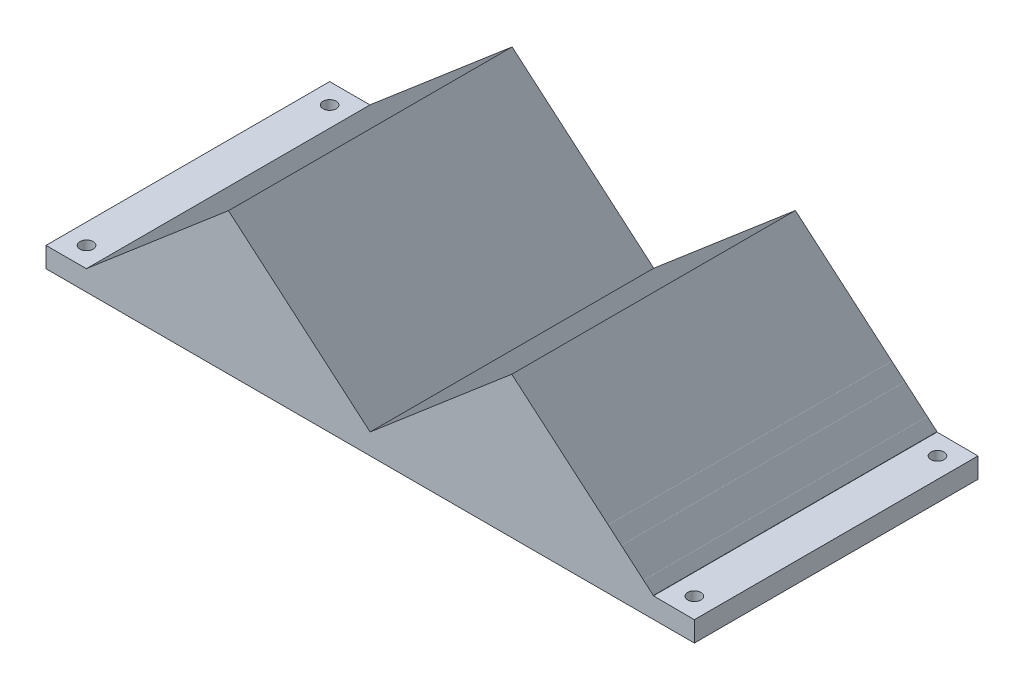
SolidWorks part; units mm, degrees
ref_plane "Front Plane" through (0, 0, 0) normal (0, 0, 1) x (1, 0, 0)
ref_plane "Top Plane" through (0, 0, 0) normal (0, 1, 0) x (1, 0, 0)
ref_plane "Right Plane" through (0, 0, 0) normal (1, 0, 0) x (0, 0, -1)
sketch "Model" plane through (0, 0, 0) normal (0, 0, 1) x (1, 0, 0)
  line L0 (0.1469, 0.2246) -> (0.2468, 0.3098)
  line L1 (0.2468, 0.3098) -> (0.3466, 0.395)
  line L2 (0.3466, 0.395) -> (0.4465, 0.4802)
  line L3 (0.4465, 0.4802) -> (0.5464, 0.5654)
  line L4 (0.5464, 0.5654) -> (0.6462, 0.6506)
  line L5 (0.6462, 0.6506) -> (0.7461, 0.7358)
  line L6 (0.7461, 0.7358) -> (0.846, 0.8209)
  line L7 (0.846, 0.8209) -> (0.9459, 0.9061)
  line L8 (0.9459, 0.9061) -> (1.0457, 0.9913)
  line L9 (1.0457, 0.9913) -> (1.1456, 1.0765)
  line L10 (1.1456, 1.0765) -> (1.2455, 1.1617)
  line L11 (1.2455, 1.1617) -> (1.3453, 1.2469)
  line L12 (1.3453, 1.2469) -> (1.4452, 1.3321)
  line L13 (1.4452, 1.3321) -> (1.5451, 1.4173)
  line L14 (1.5451, 1.4173) -> (1.645, 1.5024)
  line L15 (1.645, 1.5024) -> (1.7448, 1.5877)
  line L16 (1.7448, 1.5877) -> (1.8447, 1.6729)
  line L17 (1.8447, 1.6729) -> (1.9446, 1.758)
  line L18 (1.9446, 1.758) -> (2.0444, 1.8432)
  line L19 (2.0444, 1.8432) -> (2.1443, 1.9284)
  line L20 (2.1443, 1.9284) -> (2.2442, 2.0136)
  line L21 (2.2442, 2.0136) -> (2.3441, 2.0988)
  line L22 (2.3441, 2.0988) -> (2.4439, 2.184)
  line L23 (2.4439, 2.184) -> (2.5438, 2.2692)
  line L24 (2.5438, 2.2692) -> (2.6437, 2.3544)
  line L25 (2.6437, 2.3544) -> (2.7435, 2.4396)
  line L26 (2.7435, 2.4396) -> (2.8434, 2.5247)
  line L27 (2.8434, 2.5247) -> (2.9433, 2.61)
  line L28 (2.9433, 2.61) -> (3.0432, 2.6952)
  line L29 (3.0432, 2.6952) -> (3.143, 2.7803)
  line L30 (3.143, 2.7803) -> (3.2429, 2.8655)
  line L31 (3.2429, 2.8655) -> (3.3428, 2.9507)
  line L32 (3.3428, 2.9507) -> (3.4426, 3.0359)
  line L33 (3.4426, 3.0359) -> (3.5425, 3.1211)
  line L34 (3.5425, 3.1211) -> (3.6424, 3.2063)
  line L35 (3.6424, 3.2063) -> (3.7423, 3.2915)
  line L36 (3.7423, 3.2915) -> (3.8421, 3.3767)
  line L37 (3.8421, 3.3767) -> (3.942, 3.4619)
  line L38 (3.942, 3.4619) -> (4.0419, 3.547)
  line L39 (4.0419, 3.547) -> (4.1417, 3.6323)
  line L40 (4.1417, 3.6323) -> (4.2416, 3.7175)
  line L41 (4.2416, 3.7175) -> (4.3415, 3.8026)
  line L42 (4.3415, 3.8026) -> (4.4414, 3.8878)
  line L43 (4.4414, 3.8878) -> (4.5412, 3.973)
  line L44 (4.5412, 3.973) -> (4.6411, 4.0582)
  line L45 (4.6411, 4.0582) -> (4.741, 4.1434)
  line L46 (4.741, 4.1434) -> (4.8408, 4.2286)
  line L47 (4.8408, 4.2286) -> (4.9407, 4.3138)
  line L48 (4.9407, 4.3138) -> (5.0406, 4.399)
  line L49 (5.0406, 4.399) -> (5.1405, 4.4842)
  line L50 (5.1405, 4.4842) -> (5.2403, 4.5693)
  line L51 (5.2403, 4.5693) -> (5.3402, 4.6546)
  line L52 (5.3402, 4.6546) -> (5.4401, 4.7397)
  line L53 (5.4401, 4.7397) -> (5.5399, 4.8249)
  line L54 (5.5399, 4.8249) -> (5.6398, 4.9101)
  line L55 (5.6398, 4.9101) -> (5.7397, 4.9953)
  line L56 (5.7397, 4.9953) -> (5.8396, 5.0805)
  line L57 (5.8396, 5.0805) -> (5.9394, 5.1657)
  line L58 (5.9394, 5.1657) -> (6.0393, 5.2509)
  line L59 (6.0393, 5.2509) -> (6.1392, 5.3361)
  line L60 (6.1392, 5.3361) -> (6.239, 5.4213)
  line L61 (6.239, 5.4213) -> (6.3389, 5.5065)
  line L62 (6.3389, 5.5065) -> (6.4388, 5.5916)
  line L63 (6.4388, 5.5916) -> (6.5387, 5.6769)
  line L64 (6.5387, 5.6769) -> (6.6385, 5.762)
  line L65 (6.6385, 5.762) -> (6.7384, 5.8472)
  line L66 (6.7384, 5.8472) -> (6.8383, 5.9324)
  line L67 (6.8383, 5.9324) -> (6.9381, 6.0176)
  line L68 (6.9381, 6.0176) -> (7.038, 6.1028)
  line L69 (7.038, 6.1028) -> (7.1379, 6.188)
  line L70 (7.1379, 6.188) -> (7.2378, 6.2732)
  line L71 (7.2378, 6.2732) -> (7.3376, 6.3584)
  line L72 (7.3376, 6.3584) -> (7.4375, 6.4436)
  line L73 (7.4375, 6.4436) -> (7.5374, 6.5287)
  line L74 (7.5374, 6.5287) -> (7.6372, 6.6139)
  line L75 (7.6372, 6.6139) -> (7.7371, 6.6991)
  line L76 (7.7371, 6.6991) -> (7.837, 6.7843)
  line L77 (7.837, 6.7843) -> (7.9369, 6.8695)
  line L78 (7.9369, 6.8695) -> (8.0367, 6.9547)
  line L79 (8.0367, 6.9547) -> (8.1366, 7.0399)
  line L80 (8.1366, 7.0399) -> (8.2365, 7.1251)
  line L81 (8.2365, 7.1251) -> (8.3363, 7.2103)
  line L82 (8.3363, 7.2103) -> (8.4362, 7.2955)
  line L83 (8.4362, 7.2955) -> (8.5361, 7.3807)
  line L84 (8.5361, 7.3807) -> (8.636, 7.4659)
  line L85 (8.636, 7.4659) -> (8.7358, 7.551)
  line L86 (8.7358, 7.551) -> (8.8357, 7.6362)
  line L87 (8.8357, 7.6362) -> (8.9356, 7.7214)
  line L88 (8.9356, 7.7214) -> (9.0354, 7.8066)
  line L89 (9.0354, 7.8066) -> (9.1353, 7.8918)
  line L90 (9.1353, 7.8918) -> (9.2352, 7.977)
  line L91 (9.2352, 7.977) -> (9.3351, 8.0622)
  line L92 (9.3351, 8.0622) -> (9.4349, 8.1474)
  line L93 (9.4349, 8.1474) -> (9.5348, 8.2326)
  line L94 (9.5348, 8.2326) -> (9.6347, 8.3178)
  line L95 (9.6347, 8.3178) -> (9.7345, 8.403)
  line L96 (9.7345, 8.403) -> (9.8344, 8.4881)
  line L97 (9.8344, 8.4881) -> (9.9343, 8.5733)
  line L98 (9.9343, 8.5733) -> (10.0342, 8.6585)
  line L99 (10.0342, 8.6585) -> (10.134, 8.7437)
  line L100 (10.134, 8.7437) -> (10.2339, 8.8289)
  line L101 (10.2339, 8.8289) -> (10.3338, 8.9141)
  line L102 (10.3338, 8.9141) -> (10.4336, 8.9993)
  line L103 (10.4336, 8.9993) -> (10.5335, 9.0845)
  line L104 (10.5335, 9.0845) -> (10.6334, 9.1697)
  line L105 (10.6334, 9.1697) -> (10.7332, 9.2549)
  line L106 (10.7332, 9.2549) -> (10.8331, 9.3401)
  line L107 (10.8331, 9.3401) -> (10.933, 9.4253)
  line L108 (10.933, 9.4253) -> (11.0329, 9.5104)
  line L109 (11.0329, 9.5104) -> (11.1327, 9.5956)
  line L110 (11.1327, 9.5956) -> (11.2326, 9.6808)
  line L111 (11.2326, 9.6808) -> (11.3325, 9.766)
  line L112 (11.3325, 9.766) -> (11.4323, 9.8512)
  line L113 (11.4323, 9.8512) -> (11.5322, 9.9364)
  line L114 (11.5322, 9.9364) -> (11.6321, 10.0216)
  line L115 (11.6321, 10.0216) -> (11.732, 10.1068)
  line L116 (11.732, 10.1068) -> (11.8318, 10.192)
  line L117 (11.8318, 10.192) -> (11.9317, 10.2772)
  line L118 (11.9317, 10.2772) -> (12.0316, 10.3624)
  line L119 (12.0316, 10.3624) -> (12.1314, 10.4476)
  line L120 (12.1314, 10.4476) -> (12.2313, 10.5327)
  line L121 (12.2313, 10.5327) -> (12.3312, 10.6179)
  line L122 (12.3312, 10.6179) -> (12.4311, 10.7031)
  line L123 (12.4311, 10.7031) -> (12.5309, 10.7883)
  line L124 (12.5309, 10.7883) -> (12.6308, 10.8735)
  line L125 (12.6308, 10.8735) -> (12.7307, 10.9587)
  line L126 (12.7307, 10.9587) -> (12.8305, 11.0439)
  line L127 (12.8305, 11.0439) -> (12.9304, 11.1291)
  line L128 (12.9304, 11.1291) -> (13.0303, 11.2143)
  line L129 (13.0303, 11.2143) -> (13.1302, 11.2995)
  line L130 (13.1302, 11.2995) -> (13.23, 11.3847)
  line L131 (13.23, 11.3847) -> (13.3299, 11.4698)
  line L132 (13.3299, 11.4698) -> (13.4298, 11.555)
  line L133 (13.4298, 11.555) -> (13.5296, 11.6402)
  line L134 (13.5296, 11.6402) -> (13.6295, 11.7254)
  line L135 (13.6295, 11.7254) -> (13.7294, 11.8106)
  line L136 (13.7294, 11.8106) -> (13.8293, 11.8958)
  line L137 (13.8293, 11.8958) -> (13.9291, 11.981)
  line L138 (13.9291, 11.981) -> (14.029, 12.0662)
  line L139 (14.029, 12.0662) -> (14.1289, 12.1514)
  line L140 (14.1289, 12.1514) -> (14.2287, 12.2366)
  line L141 (14.2287, 12.2366) -> (14.3286, 12.3218)
  line L142 (14.3286, 12.3218) -> (14.4285, 12.407)
  line L143 (14.4285, 12.407) -> (14.5284, 12.4921)
  line L144 (14.5284, 12.4921) -> (14.6282, 12.5773)
  line L145 (14.6282, 12.5773) -> (14.7281, 12.6625)
  line L146 (14.7281, 12.6625) -> (14.828, 12.7477)
  line L147 (14.828, 12.7477) -> (14.9278, 12.8329)
  line L148 (14.9278, 12.8329) -> (15.0277, 12.9181)
  line L149 (15.0277, 12.9181) -> (15.1276, 13.0033)
  line L150 (15.1276, 13.0033) -> (15.2275, 13.0885)
  line L151 (15.2275, 13.0885) -> (15.3273, 13.1737)
  line L152 (15.3273, 13.1737) -> (15.4272, 13.2588)
  line L153 (15.4272, 13.2588) -> (15.5271, 13.3441)
  line L154 (15.5271, 13.3441) -> (15.6269, 13.4293)
  line L155 (15.6269, 13.4293) -> (15.7268, 13.5144)
  line L156 (15.7268, 13.5144) -> (15.8267, 13.5996)
  line L157 (15.8267, 13.5996) -> (15.9266, 13.6848)
  line L158 (15.9266, 13.6848) -> (16.0264, 13.77)
  line L159 (16.0264, 13.77) -> (16.1263, 13.8552)
  line L160 (16.1263, 13.8552) -> (16.2262, 13.9404)
  line L161 (16.2262, 13.9404) -> (16.326, 14.0256)
  line L162 (16.326, 14.0256) -> (16.4259, 14.1108)
  line L163 (16.4259, 14.1108) -> (16.5258, 14.196)
  line L164 (16.5258, 14.196) -> (16.6257, 14.2811)
  line L165 (16.6257, 14.2811) -> (16.7255, 14.3664)
  line L166 (16.7255, 14.3664) -> (16.8254, 14.4515)
  line L167 (16.8254, 14.4515) -> (16.9253, 14.5367)
  line L168 (16.9253, 14.5367) -> (17.0251, 14.6219)
  line L169 (17.0251, 14.6219) -> (17.125, 14.7071)
  line L170 (17.125, 14.7071) -> (17.2249, 14.7923)
  line L171 (17.2249, 14.7923) -> (17.3248, 14.8775)
  line L172 (17.3248, 14.8775) -> (17.4246, 14.9627)
  line L173 (17.4246, 14.9627) -> (17.5245, 15.0479)
  line L174 (17.5245, 15.0479) -> (17.6244, 15.1331)
  line L175 (17.6244, 15.1331) -> (17.7242, 15.2183)
  line L176 (17.7242, 15.2183) -> (17.8241, 15.3034)
  line L177 (17.8241, 15.3034) -> (17.924, 15.3887)
  line L178 (17.924, 15.3887) -> (18.0239, 15.4738)
  line L179 (18.0239, 15.4738) -> (18.1237, 15.559)
  line L180 (18.1237, 15.559) -> (18.2236, 15.6442)
  line L181 (18.2236, 15.6442) -> (18.3235, 15.7294)
  line L182 (18.3235, 15.7294) -> (18.4233, 15.8146)
  line L183 (18.4233, 15.8146) -> (18.5232, 15.8998)
  line L184 (18.5232, 15.8998) -> (18.6231, 15.985)
  line L185 (18.6231, 15.985) -> (18.723, 16.0702)
  line L186 (18.723, 16.0702) -> (18.8228, 16.1554)
  line L187 (18.8228, 16.1554) -> (18.9227, 16.2405)
  line L188 (18.9227, 16.2405) -> (19.0226, 16.3257)
  line L189 (19.0226, 16.3257) -> (19.1224, 16.4109)
  line L190 (19.1224, 16.4109) -> (19.2223, 16.4961)
  line L191 (19.2223, 16.4961) -> (19.3222, 16.5813)
  line L192 (19.3222, 16.5813) -> (19.422, 16.6665)
  line L193 (19.422, 16.6665) -> (19.5219, 16.7517)
  line L194 (19.5219, 16.7517) -> (19.6218, 16.8369)
  line L195 (19.6218, 16.8369) -> (19.7217, 16.9221)
  line L196 (19.7217, 16.9221) -> (19.8215, 17.0073)
  line L197 (19.8215, 17.0073) -> (19.9214, 17.0925)
  line L198 (19.9214, 17.0925) -> (20.0213, 17.1777)
  line L199 (20.0213, 17.1777) -> (20.1211, 17.2628)
  line L200 (20.1211, 17.2628) -> (20.221, 17.348)
  line L201 (20.221, 17.348) -> (20.3209, 17.4332)
  line L202 (20.3209, 17.4332) -> (20.4208, 17.5184)
  line L203 (20.4208, 17.5184) -> (20.5206, 17.6036)
  line L204 (20.5206, 17.6036) -> (20.6205, 17.6888)
  line L205 (20.6205, 17.6888) -> (20.7204, 17.774)
  line L206 (20.7204, 17.774) -> (20.8202, 17.8592)
  line L207 (20.8202, 17.8592) -> (20.9201, 17.9444)
  line L208 (20.9201, 17.9444) -> (21.02, 18.0296)
  line L209 (21.02, 18.0296) -> (21.1199, 18.1148)
  line L210 (21.1199, 18.1148) -> (21.2197, 18.2)
  line L211 (21.2197, 18.2) -> (21.3196, 18.2851)
  line L212 (21.3196, 18.2851) -> (21.4195, 18.3703)
  line L213 (21.4195, 18.3703) -> (21.5193, 18.4555)
  line L214 (21.5193, 18.4555) -> (21.6192, 18.5407)
  line L215 (21.6192, 18.5407) -> (21.7191, 18.6259)
  line L216 (21.7191, 18.6259) -> (21.819, 18.7111)
  line L217 (21.819, 18.7111) -> (21.9188, 18.7963)
  line L218 (21.9188, 18.7963) -> (22.0187, 18.8815)
  line L219 (22.0187, 18.8815) -> (22.1186, 18.9667)
  line L220 (22.1186, 18.9667) -> (22.2184, 19.0519)
  line L221 (22.2184, 19.0519) -> (22.3183, 19.1371)
  line L222 (22.3183, 19.1371) -> (22.4182, 19.2222)
  line L223 (22.4182, 19.2222) -> (22.5181, 19.3074)
  line L224 (22.5181, 19.3074) -> (22.6179, 19.3926)
  line L225 (22.6179, 19.3926) -> (22.7178, 19.4778)
  line L226 (22.7178, 19.4778) -> (22.8177, 19.563)
  line L227 (22.8177, 19.563) -> (22.9175, 19.6482)
  line L228 (22.9175, 19.6482) -> (23.0174, 19.7334)
  line L229 (23.0174, 19.7334) -> (23.1173, 19.8186)
  line L230 (23.1173, 19.8186) -> (23.2172, 19.9038)
  line L231 (23.2172, 19.9038) -> (23.317, 19.989)
  line L232 (23.317, 19.989) -> (23.4169, 20.0742)
  line L233 (23.4169, 20.0742) -> (23.5168, 20.1594)
  line L234 (23.5168, 20.1594) -> (23.6166, 20.2445)
  line L235 (23.6166, 20.2445) -> (23.7165, 20.3297)
  line L236 (23.7165, 20.3297) -> (23.8164, 20.4149)
  line L237 (23.8164, 20.4149) -> (23.9163, 20.5001)
  line L238 (23.9163, 20.5001) -> (24.0161, 20.5853)
  line L239 (24.0161, 20.5853) -> (24.116, 20.6705)
  line L240 (24.116, 20.6705) -> (24.2159, 20.7557)
  line L241 (24.2159, 20.7557) -> (24.3157, 20.8409)
  line L242 (24.3157, 20.8409) -> (24.4156, 20.9261)
  line L243 (24.4156, 20.9261) -> (24.5155, 21.0113)
  line L244 (24.5155, 21.0113) -> (24.6154, 21.0965)
  line L245 (24.6154, 21.0965) -> (24.7152, 21.1817)
  line L246 (24.7152, 21.1817) -> (24.8151, 21.2668)
  line L247 (24.8151, 21.2668) -> (24.915, 21.352)
  line L248 (24.915, 21.352) -> (25.0148, 21.4372)
  line L249 (25.0148, 21.4372) -> (25.1147, 21.5224)
  line L250 (25.1147, 21.5224) -> (25.2146, 21.6076)
  line L251 (25.2146, 21.6076) -> (25.3145, 21.6928)
  line L252 (25.3145, 21.6928) -> (25.4143, 21.778)
  line L253 (25.4143, 21.778) -> (25.5142, 21.8632)
  line L254 (25.5142, 21.8632) -> (25.6141, 21.9484)
  line L255 (25.6141, 21.9484) -> (25.7139, 22.0336)
  line L256 (25.7139, 22.0336) -> (25.8138, 22.1188)
  line L257 (25.8138, 22.1188) -> (25.9137, 22.2039)
  line L258 (25.9137, 22.2039) -> (26.0136, 22.2891)
  line L259 (26.0136, 22.2891) -> (26.1134, 22.3743)
  line L260 (26.1134, 22.3743) -> (26.2133, 22.4595)
  line L261 (26.2133, 22.4595) -> (26.3132, 22.5447)
  line L262 (26.3132, 22.5447) -> (26.413, 22.6299)
  line L263 (26.413, 22.6299) -> (26.5129, 22.7151)
  line L264 (26.5129, 22.7151) -> (26.6128, 22.8003)
  line L265 (26.6128, 22.8003) -> (26.7127, 22.8855)
  line L266 (26.7127, 22.8855) -> (26.8125, 22.9707)
  line L267 (26.8125, 22.9707) -> (26.9124, 23.0559)
  line L268 (26.9124, 23.0559) -> (27.0123, 23.1411)
  line L269 (27.0123, 23.1411) -> (27.1121, 23.2262)
  line L270 (27.1121, 23.2262) -> (27.212, 23.3114)
  line L271 (27.212, 23.3114) -> (27.3119, 23.3966)
  line L272 (27.3119, 23.3966) -> (27.4118, 23.4818)
  line L273 (27.4118, 23.4818) -> (27.5116, 23.567)
  line L274 (27.5116, 23.567) -> (27.6115, 23.6522)
  line L275 (27.6115, 23.6522) -> (27.7114, 23.7374)
  line L276 (27.7114, 23.7374) -> (27.8112, 23.8226)
  line L277 (27.8112, 23.8226) -> (27.9111, 23.9078)
  line L278 (27.9111, 23.9078) -> (28.011, 23.9929)
  line L279 (28.011, 23.9929) -> (28.1108, 24.0782)
  line L280 (28.1108, 24.0782) -> (28.2107, 24.1634)
  line L281 (28.2107, 24.1634) -> (28.3106, 24.2485)
  line L282 (28.3106, 24.2485) -> (28.4105, 24.3337)
  line L283 (28.4105, 24.3337) -> (28.5103, 24.4189)
  line L284 (28.5103, 24.4189) -> (28.6102, 24.5041)
  line L285 (28.6102, 24.5041) -> (28.7101, 24.5893)
  line L286 (28.7101, 24.5893) -> (28.8099, 24.6745)
  line L287 (28.8099, 24.6745) -> (28.9098, 24.7597)
  line L288 (28.9098, 24.7597) -> (29.0097, 24.8449)
  line L289 (29.0097, 24.8449) -> (29.1096, 24.9301)
  line L290 (29.1096, 24.9301) -> (29.2094, 25.0152)
  line L291 (29.2094, 25.0152) -> (29.3093, 25.1005)
  line L292 (29.3093, 25.1005) -> (29.4092, 25.1856)
  line L293 (29.4092, 25.1856) -> (29.509, 25.2708)
  line L294 (29.509, 25.2708) -> (29.6089, 25.356)
  line L295 (29.6089, 25.356) -> (29.7088, 25.4412)
  line L296 (29.7088, 25.4412) -> (29.8087, 25.5264)
  line L297 (29.8087, 25.5264) -> (29.9085, 25.6116)
  line L298 (29.9085, 25.6116) -> (30.0084, 25.6968)
  line L299 (30.0084, 25.6968) -> (30.1083, 25.782)
  line L300 (30.1083, 25.782) -> (30.2081, 25.8672)
  line L301 (30.2081, 25.8672) -> (30.308, 25.9524)
  line L302 (30.308, 25.9524) -> (30.4079, 26.0375)
  line L303 (30.4079, 26.0375) -> (30.5078, 26.1228)
  line L304 (30.5078, 26.1228) -> (30.6076, 26.2079)
  line L305 (30.6076, 26.2079) -> (30.7075, 26.2931)
  line L306 (30.7075, 26.2931) -> (30.8074, 26.3783)
  line L307 (30.8074, 26.3783) -> (30.9072, 26.4635)
  line L308 (30.9072, 26.4635) -> (31.0071, 26.5487)
  line L309 (31.0071, 26.5487) -> (31.107, 26.6339)
  line L310 (31.107, 26.6339) -> (31.2069, 26.7191)
  line L311 (31.2069, 26.7191) -> (31.3067, 26.8043)
  line L312 (31.3067, 26.8043) -> (31.4066, 26.8895)
  line L313 (31.4066, 26.8895) -> (31.5065, 26.9746)
  line L314 (31.5065, 26.9746) -> (31.6063, 27.0598)
  line L315 (31.6063, 27.0598) -> (31.7062, 27.1451)
  line L316 (31.7062, 27.1451) -> (31.8061, 27.2302)
  line L317 (31.8061, 27.2302) -> (31.906, 27.3154)
  line L318 (31.906, 27.3154) -> (32.0058, 27.4006)
  line L319 (32.0058, 27.4006) -> (32.1057, 27.4858)
  line L320 (32.1057, 27.4858) -> (32.2056, 27.571)
  line L321 (32.2056, 27.571) -> (32.3054, 27.6562)
  line L322 (32.3054, 27.6562) -> (32.4053, 27.7414)
  line L323 (32.4053, 27.7414) -> (32.5052, 27.8266)
  line L324 (32.5052, 27.8266) -> (32.6051, 27.9118)
  line L325 (32.6051, 27.9118) -> (32.7049, 27.9969)
  line L326 (32.7049, 27.9969) -> (32.8048, 28.0821)
  line L327 (32.8048, 28.0821) -> (32.9047, 28.1673)
  line L328 (32.9047, 28.1673) -> (33.0045, 28.2525)
  line L329 (33.0045, 28.2525) -> (33.1044, 28.3377)
  line L330 (33.1044, 28.3377) -> (33.2043, 28.4229)
  line L331 (33.2043, 28.4229) -> (33.3042, 28.5081)
  line L332 (33.3042, 28.5081) -> (33.404, 28.5933)
  line L333 (33.404, 28.5933) -> (33.5039, 28.6785)
  line L334 (33.5039, 28.6785) -> (33.6038, 28.7637)
  line L335 (33.6038, 28.7637) -> (33.7036, 28.8489)
  line L336 (33.7036, 28.8489) -> (33.8035, 28.9341)
  line L337 (33.8035, 28.9341) -> (33.9034, 29.0192)
  line L338 (33.9034, 29.0192) -> (34.0033, 29.1044)
  line L339 (34.0033, 29.1044) -> (34.1031, 29.1896)
  line L340 (34.1031, 29.1896) -> (34.203, 29.2748)
  line L341 (34.203, 29.2748) -> (34.3029, 29.36)
  line L342 (34.3029, 29.36) -> (34.4027, 29.4452)
  line L343 (34.4027, 29.4452) -> (34.5026, 29.5304)
  line L344 (34.5026, 29.5304) -> (34.6025, 29.6156)
  line L345 (34.6025, 29.6156) -> (34.7024, 29.7008)
  line L346 (34.7024, 29.7008) -> (34.8022, 29.786)
  line L347 (34.8022, 29.786) -> (34.9021, 29.8712)
  line L348 (34.9021, 29.8712) -> (35.002, 29.9563)
  line L349 (35.002, 29.9563) -> (35.1018, 30.0415)
  line L350 (35.1018, 30.0415) -> (35.2017, 30.1267)
  line L351 (35.2017, 30.1267) -> (35.3016, 30.2119)
  line L352 (35.3016, 30.2119) -> (35.4015, 30.2971)
  line L353 (35.4015, 30.2971) -> (35.5013, 30.3823)
  line L354 (35.5013, 30.3823) -> (35.6012, 30.4675)
  line L355 (35.6012, 30.4675) -> (35.7011, 30.5527)
  line L356 (35.7011, 30.5527) -> (35.8009, 30.6379)
  line L357 (35.8009, 30.6379) -> (35.9008, 30.7231)
  line L358 (35.9008, 30.7231) -> (36.0007, 30.8083)
  line L359 (36.0007, 30.8083) -> (36.1006, 30.8935)
  line L360 (36.1006, 30.8935) -> (36.2004, 30.9786)
  line L361 (36.2004, 30.9786) -> (36.3003, 31.0638)
  line L362 (36.3003, 31.0638) -> (36.4002, 31.149)
  line L363 (36.4002, 31.149) -> (36.5, 31.2342)
  line L364 (36.5, 31.2342) -> (36.5999, 31.3194)
  line L365 (36.5999, 31.3194) -> (36.6998, 31.4046)
  line L366 (36.6998, 31.4046) -> (36.7996, 31.4898)
  line L367 (36.7996, 31.4898) -> (36.8995, 31.575)
  line L368 (36.8995, 31.575) -> (36.9994, 31.6602)
  line L369 (36.9994, 31.6602) -> (37.0993, 31.7453)
  line L370 (37.0993, 31.7453) -> (37.1991, 31.8306)
  line L371 (37.1991, 31.8306) -> (37.299, 31.9158)
  line L372 (37.299, 31.9158) -> (37.3989, 32.0009)
  line L373 (37.3989, 32.0009) -> (37.4987, 32.0861)
  line L374 (37.4987, 32.0861) -> (37.5986, 32.1713)
  line L375 (37.5986, 32.1713) -> (37.6985, 32.2565)
  line L376 (37.6985, 32.2565) -> (37.7984, 32.3417)
  line L377 (37.7984, 32.3417) -> (37.8982, 32.4269)
  line L378 (37.8982, 32.4269) -> (37.9981, 32.5121)
  line L379 (37.9981, 32.5121) -> (38.098, 32.5973)
  line L380 (38.098, 32.5973) -> (38.1978, 32.6825)
  line L381 (38.1978, 32.6825) -> (38.2977, 32.7677)
  line L382 (38.2977, 32.7677) -> (38.3976, 32.8529)
  line L383 (38.3976, 32.8529) -> (38.4975, 32.938)
  line L384 (38.4975, 32.938) -> (38.5973, 33.0232)
  line L385 (38.5973, 33.0232) -> (38.6972, 33.1084)
  line L386 (38.6972, 33.1084) -> (38.7971, 33.1936)
  line L387 (38.7971, 33.1936) -> (38.8969, 33.2788)
  line L388 (38.8969, 33.2788) -> (38.9968, 33.364)
  line L389 (38.9968, 33.364) -> (39.0967, 33.4492)
  line L390 (39.0967, 33.4492) -> (39.1966, 33.5344)
  line L391 (39.1966, 33.5344) -> (39.2964, 33.6196)
  line L392 (39.2964, 33.6196) -> (39.3963, 33.7048)
  line L393 (39.3963, 33.7048) -> (39.4962, 33.7899)
  line L394 (39.4962, 33.7899) -> (39.596, 33.8752)
  line L395 (39.596, 33.8752) -> (39.6959, 33.9603)
  line L396 (39.6959, 33.9603) -> (39.7958, 34.0455)
  line L397 (39.7958, 34.0455) -> (39.8957, 34.1307)
  line L398 (39.8957, 34.1307) -> (39.9955, 34.2159)
  line L399 (39.9955, 34.2159) -> (40.0954, 34.3011)
  line L400 (40.0954, 34.3011) -> (40.1953, 34.3863)
  line L401 (40.1953, 34.3863) -> (40.2951, 34.4715)
  line L402 (40.2951, 34.4715) -> (40.395, 34.5567)
  line L403 (40.395, 34.5567) -> (40.4949, 34.6419)
  line L404 (40.4949, 34.6419) -> (40.5948, 34.7271)
  line L405 (40.5948, 34.7271) -> (40.6946, 34.8123)
  line L406 (40.6946, 34.8123) -> (40.7945, 34.8975)
  line L407 (40.7945, 34.8975) -> (40.8944, 34.9826)
  line L408 (40.8944, 34.9826) -> (40.9942, 35.0678)
  line L409 (40.9942, 35.0678) -> (41.0941, 35.153)
  line L410 (41.0941, 35.153) -> (41.194, 35.2382)
  line L411 (41.194, 35.2382) -> (41.2939, 35.3234)
  line L412 (41.2939, 35.3234) -> (41.3937, 35.4086)
  line L413 (41.3937, 35.4086) -> (41.4936, 35.4938)
  line L414 (41.4936, 35.4938) -> (41.5935, 35.579)
  line L415 (41.5935, 35.579) -> (41.6933, 35.6642)
  line L416 (41.6933, 35.6642) -> (41.7932, 35.7493)
  line L417 (41.7932, 35.7493) -> (41.8931, 35.8346)
  line L418 (41.8931, 35.8346) -> (41.993, 35.9197)
  line L419 (41.993, 35.9197) -> (42.0928, 36.0049)
  line L420 (42.0928, 36.0049) -> (42.1927, 36.0901)
  line L421 (42.1927, 36.0901) -> (42.2926, 36.1753)
  line L422 (42.2926, 36.1753) -> (42.3924, 36.2605)
  line L423 (42.3924, 36.2605) -> (42.4923, 36.3457)
  line L424 (42.4923, 36.3457) -> (42.5922, 36.4309)
  line L425 (42.5922, 36.4309) -> (42.6921, 36.5161)
  line L426 (42.6921, 36.5161) -> (42.7919, 36.6013)
  line L427 (42.7919, 36.6013) -> (42.8918, 36.6865)
  line L428 (42.8918, 36.6865) -> (42.9917, 36.7716)
  line L429 (42.9917, 36.7716) -> (43.0915, 36.8569)
  line L430 (43.0915, 36.8569) -> (43.1914, 36.942)
  line L431 (43.1914, 36.942) -> (43.2913, 37.0272)
  line L432 (43.2913, 37.0272) -> (43.3912, 37.1124)
  line L433 (43.3912, 37.1124) -> (43.491, 37.1976)
  line L434 (43.491, 37.1976) -> (43.5909, 37.2828)
  line L435 (43.5909, 37.2828) -> (43.6908, 37.368)
  line L436 (43.6908, 37.368) -> (43.7906, 37.4532)
  line L437 (43.7906, 37.4532) -> (43.8905, 37.5384)
  line L438 (43.8905, 37.5384) -> (43.9904, 37.6236)
  line L439 (43.9904, 37.6236) -> (44.0903, 37.7087)
  line L440 (44.0903, 37.7087) -> (44.1901, 37.7939)
  line L441 (44.1901, 37.7939) -> (44.29, 37.8792)
  line L442 (44.29, 37.8792) -> (44.3899, 37.9643)
  line L443 (44.3899, 37.9643) -> (44.4897, 38.0495)
  line L444 (44.4897, 38.0495) -> (44.5896, 38.1347)
  line L445 (44.5896, 38.1347) -> (44.6895, 38.2199)
  line L446 (44.6895, 38.2199) -> (44.7894, 38.3051)
  line L447 (44.7894, 38.3051) -> (44.8892, 38.3903)
  line L448 (44.8892, 38.3903) -> (44.9891, 38.4755)
  line L449 (44.9891, 38.4755) -> (45.089, 38.5607)
  line L450 (45.089, 38.5607) -> (45.1888, 38.6459)
  line L451 (45.1888, 38.6459) -> (45.2887, 38.731)
  line L452 (45.2887, 38.731) -> (45.3886, 38.8162)
  line L453 (45.3886, 38.8162) -> (45.4885, 38.9014)
  line L454 (45.4885, 38.9014) -> (45.5883, 38.9866)
  line L455 (45.5883, 38.9866) -> (45.6882, 39.0718)
  line L456 (45.6882, 39.0718) -> (45.7881, 39.157)
  line L457 (45.7881, 39.157) -> (45.8879, 39.2422)
  line L458 (45.8879, 39.2422) -> (45.9878, 39.3274)
  line L459 (45.9878, 39.3274) -> (46.0877, 39.4126)
  line L460 (46.0877, 39.4126) -> (46.1875, 39.4978)
  line L461 (46.1875, 39.4978) -> (46.2874, 39.583)
  line L462 (46.2874, 39.583) -> (46.3873, 39.6682)
  line L463 (46.3873, 39.6682) -> (46.4872, 39.7533)
  line L464 (46.4872, 39.7533) -> (46.587, 39.8385)
  line L465 (46.587, 39.8385) -> (46.6869, 39.9237)
  line L466 (46.6869, 39.9237) -> (46.7868, 40.0089)
  line L467 (46.7868, 40.0089) -> (46.8866, 40.0941)
  line L468 (46.8866, 40.0941) -> (46.9865, 40.1793)
  line L469 (46.9865, 40.1793) -> (47.0864, 40.2645)
  line L470 (47.0864, 40.2645) -> (47.1863, 40.3497)
  line L471 (47.1863, 40.3497) -> (47.2861, 40.4349)
  line L472 (47.2861, 40.4349) -> (47.386, 40.5201)
  line L473 (47.386, 40.5201) -> (47.4859, 40.6053)
  line L474 (47.4859, 40.6053) -> (47.5857, 40.6904)
  line L475 (47.5857, 40.6904) -> (47.6856, 40.7756)
  line L476 (47.6856, 40.7756) -> (47.7855, 40.8608)
  line L477 (47.7855, 40.8608) -> (47.8854, 40.946)
  line L478 (47.8854, 40.946) -> (47.9852, 41.0312)
  line L479 (47.9852, 41.0312) -> (48.0851, 41.1164)
  line L480 (48.0851, 41.1164) -> (48.185, 41.2016)
  line L481 (48.185, 41.2016) -> (48.2848, 41.2868)
  line L482 (48.2848, 41.2868) -> (48.3847, 41.372)
  line L483 (48.3847, 41.372) -> (48.4846, 41.4572)
  line L484 (48.4846, 41.4572) -> (48.5845, 41.5424)
  line L485 (48.5845, 41.5424) -> (48.6843, 41.6276)
  line L486 (48.6843, 41.6276) -> (48.7842, 41.7127)
  line L487 (48.7842, 41.7127) -> (48.8841, 41.7979)
  line L488 (48.8841, 41.7979) -> (48.9839, 41.8831)
  line L489 (48.9839, 41.8831) -> (49.0838, 41.9683)
  line L490 (49.0838, 41.9683) -> (49.1837, 42.0535)
  line L491 (49.1837, 42.0535) -> (49.2836, 42.1387)
  line L492 (49.2836, 42.1387) -> (49.3834, 42.2239)
  line L493 (49.3834, 42.2239) -> (49.4833, 42.3091)
  line L494 (49.4833, 42.3091) -> (49.5832, 42.3943)
  line L495 (49.5832, 42.3943) -> (49.683, 42.4794)
  line L496 (49.683, 42.4794) -> (49.7829, 42.5647)
  line L497 (49.7829, 42.5647) -> (49.8828, 42.6499)
  line L498 (49.8828, 42.6499) -> (49.9827, 42.735)
  line L499 (49.9827, 42.735) -> (50.0825, 42.8202)
  line L500 (50.0825, 42.8202) -> (50.1824, 42.9054)
  line L501 (50.1824, 42.9054) -> (50.2823, 42.9906)
  line L502 (50.2823, 42.9906) -> (50.3821, 43.0758)
  line L503 (50.3821, 43.0758) -> (50.482, 43.161)
  line L504 (50.482, 43.161) -> (50.5819, 43.2462)
  line L505 (50.5819, 43.2462) -> (50.6818, 43.3314)
  line L506 (50.6818, 43.3314) -> (50.7816, 43.4166)
  line L507 (50.7816, 43.4166) -> (50.8815, 43.5017)
  line L508 (50.8815, 43.5017) -> (50.9814, 43.587)
  line L509 (50.9814, 43.587) -> (51.0812, 43.6721)
  line L510 (51.0812, 43.6721) -> (51.1811, 43.7573)
  line L511 (51.1811, 43.7573) -> (51.281, 43.8425)
  line L512 (51.281, 43.8425) -> (51.3809, 43.9277)
  line L513 (51.3809, 43.9277) -> (51.4807, 44.0129)
  line L514 (51.4807, 44.0129) -> (51.5806, 44.0981)
  line L515 (51.5806, 44.0981) -> (51.6805, 44.1833)
  line L516 (51.6805, 44.1833) -> (51.7803, 44.2685)
  line L517 (51.7803, 44.2685) -> (51.8802, 44.3537)
  line L518 (51.8802, 44.3537) -> (51.9801, 44.4388)
  line L519 (51.9801, 44.4388) -> (52.08, 44.524)
  line L520 (52.08, 44.524) -> (52.1798, 44.6093)
  line L521 (52.1798, 44.6093) -> (52.2797, 44.6944)
  line L522 (52.2797, 44.6944) -> (52.3796, 44.7796)
  line L523 (52.3796, 44.7796) -> (52.4794, 44.8648)
  line L524 (52.4794, 44.8648) -> (52.5793, 44.95)
  line L525 (52.5793, 44.95) -> (52.6792, 45.0352)
  line L526 (52.6792, 45.0352) -> (52.7791, 45.1204)
  line L527 (52.7791, 45.1204) -> (52.8789, 45.2056)
  line L528 (52.8789, 45.2056) -> (52.9788, 45.2908)
  line L529 (52.9788, 45.2908) -> (53.0787, 45.376)
  line L530 (53.0787, 45.376) -> (53.1785, 45.4612)
  line L531 (53.1785, 45.4612) -> (53.2784, 45.5463)
  line L532 (53.2784, 45.5463) -> (53.3783, 45.6316)
  line L533 (53.3783, 45.6316) -> (53.4782, 45.7167)
  line L534 (53.4782, 45.7167) -> (53.578, 45.8019)
  line L535 (53.578, 45.8019) -> (53.6779, 45.8871)
  line L536 (53.6779, 45.8871) -> (53.7778, 45.9723)
  line L537 (53.7778, 45.9723) -> (53.8776, 46.0575)
  line L538 (53.8776, 46.0575) -> (53.9775, 46.1427)
  line L539 (53.9775, 46.1427) -> (54.0774, 46.2279)
  line L540 (54.0774, 46.2279) -> (54.1773, 46.3131)
  line L541 (54.1773, 46.3131) -> (54.2771, 46.3983)
  line L542 (54.2771, 46.3983) -> (54.377, 46.4834)
  line L543 (54.377, 46.4834) -> (54.4769, 46.5686)
  line L544 (54.4769, 46.5686) -> (54.5767, 46.6538)
  line L545 (54.5767, 46.6538) -> (54.6766, 46.739)
  line L546 (54.6766, 46.739) -> (54.7765, 46.8242)
  line L547 (54.7765, 46.8242) -> (54.8764, 46.9094)
  line L548 (54.8764, 46.9094) -> (54.9762, 46.9946)
  line L549 (54.9762, 46.9946) -> (55.0761, 47.0798)
  line L550 (55.0761, 47.0798) -> (55.176, 47.165)
  line L551 (55.176, 47.165) -> (55.2758, 47.2502)
  line L552 (55.2758, 47.2502) -> (55.3757, 47.3354)
  line L553 (55.3757, 47.3354) -> (55.4756, 47.4206)
  line L554 (55.4756, 47.4206) -> (55.5754, 47.5057)
  line L555 (55.5754, 47.5057) -> (55.6753, 47.5909)
  line L556 (55.6753, 47.5909) -> (55.7752, 47.6761)
  line L557 (55.7752, 47.6761) -> (55.8751, 47.7613)
  line L558 (55.8751, 47.7613) -> (55.9749, 47.8465)
  line L559 (55.9749, 47.8465) -> (56.0748, 47.9317)
  line L560 (56.0748, 47.9317) -> (56.1747, 48.0169)
  line L561 (56.1747, 48.0169) -> (56.2745, 48.1021)
  line L562 (56.2745, 48.1021) -> (56.3744, 48.1873)
  line L563 (56.3744, 48.1873) -> (56.4743, 48.2725)
  line L564 (56.4743, 48.2725) -> (56.5742, 48.3577)
  line L565 (56.5742, 48.3577) -> (56.674, 48.4428)
  line L566 (56.674, 48.4428) -> (56.7739, 48.528)
  line L567 (56.7739, 48.528) -> (56.8738, 48.6132)
  line L568 (56.8738, 48.6132) -> (56.9736, 48.6984)
  line L569 (56.9736, 48.6984) -> (57.0735, 48.7836)
  line L570 (57.0735, 48.7836) -> (57.1734, 48.8688)
  line L571 (57.1734, 48.8688) -> (57.2733, 48.954)
  line L572 (57.2733, 48.954) -> (57.3731, 49.0392)
  line L573 (57.3731, 49.0392) -> (57.473, 49.1244)
  line L574 (57.473, 49.1244) -> (57.5729, 49.2096)
  line L575 (57.5729, 49.2096) -> (57.6727, 49.2948)
  line L576 (57.6727, 49.2948) -> (57.7726, 49.38)
  line L577 (57.7726, 49.38) -> (57.8725, 49.4651)
  line L578 (57.8725, 49.4651) -> (57.9724, 49.5503)
  line L579 (57.9724, 49.5503) -> (58.0722, 49.6355)
  line L580 (58.0722, 49.6355) -> (58.1721, 49.7207)
  line L581 (58.1721, 49.7207) -> (58.272, 49.8059)
  line L582 (58.272, 49.8059) -> (58.3718, 49.8911)
  line L583 (58.3718, 49.8911) -> (58.4717, 49.9763)
  line L584 (58.4717, 49.9763) -> (58.5716, 50.0615)
  line L585 (58.5716, 50.0615) -> (58.6715, 50.1467)
  line L586 (58.6715, 50.1467) -> (58.7713, 50.2319)
  line L587 (58.7713, 50.2319) -> (58.8712, 50.3171)
  line L588 (58.8712, 50.3171) -> (58.9711, 50.4023)
  line L589 (58.9711, 50.4023) -> (59.0709, 50.4874)
  line L590 (59.0709, 50.4874) -> (59.1708, 50.5726)
  line L591 (59.1708, 50.5726) -> (59.2707, 50.6578)
  line L592 (59.2707, 50.6578) -> (59.3706, 50.743)
  line L593 (59.3706, 50.743) -> (59.4704, 50.8282)
  line L594 (59.4704, 50.8282) -> (59.5703, 50.9134)
  line L595 (59.5703, 50.9134) -> (59.6702, 50.9986)
  line L596 (59.6702, 50.9986) -> (59.77, 51.0838)
  line L597 (59.77, 51.0838) -> (59.8699, 51.169)
  line L598 (59.8699, 51.169) -> (59.9698, 51.2542)
  line L599 (59.9698, 51.2542) -> (60.0697, 51.3394)
  line L600 (60.0697, 51.3394) -> (60.1695, 51.4245)
  line L601 (60.1695, 51.4245) -> (60.2694, 51.5097)
  line L602 (60.2694, 51.5097) -> (60.3693, 51.5949)
  line L603 (60.3693, 51.5949) -> (60.4691, 51.6801)
  line L604 (60.4691, 51.6801) -> (60.569, 51.7653)
  line L605 (60.569, 51.7653) -> (60.6689, 51.8505)
  line L606 (60.6689, 51.8505) -> (60.7688, 51.9357)
  line L607 (60.7688, 51.9357) -> (60.8686, 52.0209)
  line L608 (60.8686, 52.0209) -> (60.9685, 52.1061)
  line L609 (60.9685, 52.1061) -> (61.0684, 52.1913)
  line L610 (61.0684, 52.1913) -> (61.1682, 52.2765)
  line L611 (61.1682, 52.2765) -> (61.2681, 52.3617)
  line L612 (61.2681, 52.3617) -> (61.368, 52.4468)
  line L613 (61.368, 52.4468) -> (61.4679, 52.532)
  line L614 (61.4679, 52.532) -> (61.5677, 52.6172)
  line L615 (61.5677, 52.6172) -> (61.6676, 52.7024)
  line L616 (61.6676, 52.7024) -> (61.7675, 52.7876)
  line L617 (61.7675, 52.7876) -> (61.8673, 52.8728)
  line L618 (61.8673, 52.8728) -> (61.9672, 52.958)
  line L619 (61.9672, 52.958) -> (62.0671, 53.0432)
  line L620 (62.0671, 53.0432) -> (62.167, 53.1284)
  line L621 (62.167, 53.1284) -> (62.2668, 53.2135)
  line L622 (62.2668, 53.2135) -> (62.3667, 53.2988)
  line L623 (62.3667, 53.2988) -> (62.4666, 53.384)
  line L624 (62.4666, 53.384) -> (62.5664, 53.4691)
  line L625 (62.5664, 53.4691) -> (62.6663, 53.5543)
  line L626 (62.6663, 53.5543) -> (62.7662, 53.6395)
  line L627 (62.7662, 53.6395) -> (62.8661, 53.7247)
  line L628 (62.8661, 53.7247) -> (62.9659, 53.8099)
  line L629 (62.9659, 53.8099) -> (63.0658, 53.8951)
  line L630 (63.0658, 53.8951) -> (63.1657, 53.9803)
  line L631 (63.1657, 53.9803) -> (63.2655, 54.0655)
  line L632 (63.2655, 54.0655) -> (63.3654, 54.1507)
  line L633 (63.3654, 54.1507) -> (63.4653, 54.2358)
  line L634 (63.4653, 54.2358) -> (63.5652, 54.3211)
  line L635 (63.5652, 54.3211) -> (63.665, 54.4062)
  line L636 (63.665, 54.4062) -> (63.7649, 54.4914)
  line L637 (63.7649, 54.4914) -> (63.8648, 54.5766)
  line L638 (63.8648, 54.5766) -> (63.9646, 54.6618)
  line L639 (63.9646, 54.6618) -> (64.0645, 54.747)
  line L640 (64.0645, 54.747) -> (64.1644, 54.8322)
  line L641 (64.1644, 54.8322) -> (64.2642, 54.9174)
  line L642 (64.2642, 54.9174) -> (64.3641, 55.0026)
  line L643 (64.3641, 55.0026) -> (64.464, 55.0878)
  line L644 (64.464, 55.0878) -> (64.5639, 55.173)
  line L645 (64.5639, 55.173) -> (64.6637, 55.2581)
  line L646 (64.6637, 55.2581) -> (64.7636, 55.3434)
  line L647 (64.7636, 55.3434) -> (64.8635, 55.4285)
  line L648 (64.8635, 55.4285) -> (64.9633, 55.5137)
  line L649 (64.9633, 55.5137) -> (65.0632, 55.5989)
  line L650 (65.0632, 55.5989) -> (65.1631, 55.6841)
  line L651 (65.1631, 55.6841) -> (65.263, 55.7693)
  line L652 (65.263, 55.7693) -> (65.3628, 55.8545)
  line L653 (65.3628, 55.8545) -> (65.4627, 55.9397)
  line L654 (65.4627, 55.9397) -> (65.5626, 56.0249)
  line L655 (65.5626, 56.0249) -> (65.6624, 56.1101)
  line L656 (65.6624, 56.1101) -> (65.7623, 56.1952)
  line L657 (65.7623, 56.1952) -> (65.8622, 56.2804)
  line L658 (65.8622, 56.2804) -> (65.9621, 56.3657)
  line L659 (65.9621, 56.3657) -> (66.0619, 56.4508)
  line L660 (66.0619, 56.4508) -> (66.1618, 56.536)
  line L661 (66.1618, 56.536) -> (66.2617, 56.6212)
  line L662 (66.2617, 56.6212) -> (66.3615, 56.7064)
  line L663 (66.3615, 56.7064) -> (66.4614, 56.7916)
  line L664 (66.4614, 56.7916) -> (66.5613, 56.8768)
  line L665 (66.5613, 56.8768) -> (66.6612, 56.962)
  line L666 (66.6612, 56.962) -> (66.761, 57.0472)
  line L667 (66.761, 57.0472) -> (66.8609, 57.1324)
  line L668 (66.8609, 57.1324) -> (66.9608, 57.2175)
  line L669 (66.9608, 57.2175) -> (67.0606, 57.3027)
  line L670 (67.0606, 57.3027) -> (67.1605, 57.3879)
  line L671 (67.1605, 57.3879) -> (67.2604, 57.4731)
  line L672 (67.2604, 57.4731) -> (67.3603, 57.5583)
  line L673 (67.3603, 57.5583) -> (67.4601, 57.6435)
  line L674 (67.4601, 57.6435) -> (67.56, 57.7287)
  line L675 (67.56, 57.7287) -> (67.6599, 57.8139)
  line L676 (67.6599, 57.8139) -> (67.7597, 57.8991)
  line L677 (67.7597, 57.8991) -> (67.8596, 57.9843)
  line L678 (67.8596, 57.9843) -> (67.9595, 58.0695)
  line L679 (67.9595, 58.0695) -> (68.0594, 58.1547)
  line L680 (68.0594, 58.1547) -> (68.1592, 58.2398)
  line L681 (68.1592, 58.2398) -> (68.2591, 58.325)
  line L682 (68.2591, 58.325) -> (68.359, 58.4102)
  line L683 (68.359, 58.4102) -> (68.4588, 58.4954)
  line L684 (68.4588, 58.4954) -> (68.5587, 58.5806)
  line L685 (68.5587, 58.5806) -> (68.6586, 58.6658)
  line L686 (68.6586, 58.6658) -> (68.7585, 58.751)
  line L687 (68.7585, 58.751) -> (68.8583, 58.8362)
  line L688 (68.8583, 58.8362) -> (68.9582, 58.9214)
  line L689 (68.9582, 58.9214) -> (69.0581, 59.0066)
  line L690 (69.0581, 59.0066) -> (69.1579, 59.0918)
  line L691 (69.1579, 59.0918) -> (69.2578, 59.1769)
  line L692 (69.2578, 59.1769) -> (69.3577, 59.2621)
  line L693 (69.3577, 59.2621) -> (69.4576, 59.3473)
  line L694 (69.4576, 59.3473) -> (69.5574, 59.4325)
  line L695 (69.5574, 59.4325) -> (69.6573, 59.5177)
  line L696 (69.6573, 59.5177) -> (69.7572, 59.6029)
  line L697 (69.7572, 59.6029) -> (69.857, 59.6881)
  line L698 (69.857, 59.6881) -> (69.9569, 59.7733)
  line L699 (69.9569, 59.7733) -> (70.0568, 59.8585)
  line L700 (70.0568, 59.8585) -> (70.1567, 59.7733)
  line L701 (70.1567, 59.7733) -> (70.2565, 59.6881)
  line L702 (70.2565, 59.6881) -> (70.3564, 59.6029)
  line L703 (70.3564, 59.6029) -> (70.4563, 59.5177)
  line L704 (70.4563, 59.5177) -> (70.5561, 59.4325)
  line L705 (70.5561, 59.4325) -> (70.656, 59.3473)
  line L706 (70.656, 59.3473) -> (70.7559, 59.2621)
  line L707 (70.7559, 59.2621) -> (70.8558, 59.1769)
  line L708 (70.8558, 59.1769) -> (70.9556, 59.0918)
  line L709 (70.9556, 59.0918) -> (71.0555, 59.0066)
  line L710 (71.0555, 59.0066) -> (71.1554, 58.9214)
  line L711 (71.1554, 58.9214) -> (71.2552, 58.8362)
  line L712 (71.2552, 58.8362) -> (71.3551, 58.751)
  line L713 (71.3551, 58.751) -> (71.455, 58.6658)
  line L714 (71.455, 58.6658) -> (71.5549, 58.5806)
  line L715 (71.5549, 58.5806) -> (71.6547, 58.4954)
  line L716 (71.6547, 58.4954) -> (71.7546, 58.4102)
  line L717 (71.7546, 58.4102) -> (71.8545, 58.325)
  line L718 (71.8545, 58.325) -> (71.9543, 58.2398)
  line L719 (71.9543, 58.2398) -> (72.0542, 58.1547)
  line L720 (72.0542, 58.1547) -> (72.1541, 58.0695)
  line L721 (72.1541, 58.0695) -> (72.254, 57.9843)
  line L722 (72.254, 57.9843) -> (72.3538, 57.8991)
  line L723 (72.3538, 57.8991) -> (72.4537, 57.8139)
  line L724 (72.4537, 57.8139) -> (72.5536, 57.7287)
  line L725 (72.5536, 57.7287) -> (72.6534, 57.6435)
  line L726 (72.6534, 57.6435) -> (72.7533, 57.5583)
  line L727 (72.7533, 57.5583) -> (72.8532, 57.4731)
  line L728 (72.8532, 57.4731) -> (72.9531, 57.3879)
  line L729 (72.9531, 57.3879) -> (73.0529, 57.3027)
  line L730 (73.0529, 57.3027) -> (73.1528, 57.2175)
  line L731 (73.1528, 57.2175) -> (73.2527, 57.1324)
  line L732 (73.2527, 57.1324) -> (73.3525, 57.0472)
  line L733 (73.3525, 57.0472) -> (73.4524, 56.962)
  line L734 (73.4524, 56.962) -> (73.5523, 56.8768)
  line L735 (73.5523, 56.8768) -> (73.6521, 56.7916)
  line L736 (73.6521, 56.7916) -> (73.752, 56.7064)
  line L737 (73.752, 56.7064) -> (73.8519, 56.6212)
  line L738 (73.8519, 56.6212) -> (73.9518, 56.536)
  line L739 (73.9518, 56.536) -> (74.0516, 56.4508)
  line L740 (74.0516, 56.4508) -> (74.1515, 56.3657)
  line L741 (74.1515, 56.3657) -> (74.2514, 56.2804)
  line L742 (74.2514, 56.2804) -> (74.3512, 56.1952)
  line L743 (74.3512, 56.1952) -> (74.4511, 56.1101)
  line L744 (74.4511, 56.1101) -> (74.551, 56.0249)
  line L745 (74.551, 56.0249) -> (74.6509, 55.9397)
  line L746 (74.6509, 55.9397) -> (74.7507, 55.8545)
  line L747 (74.7507, 55.8545) -> (74.8506, 55.7693)
  line L748 (74.8506, 55.7693) -> (74.9505, 55.6841)
  line L749 (74.9505, 55.6841) -> (75.0503, 55.5989)
  line L750 (75.0503, 55.5989) -> (75.1502, 55.5137)
  line L751 (75.1502, 55.5137) -> (75.2501, 55.4285)
  line L752 (75.2501, 55.4285) -> (75.35, 55.3434)
  line L753 (75.35, 55.3434) -> (75.4498, 55.2581)
  line L754 (75.4498, 55.2581) -> (75.5497, 55.173)
  line L755 (75.5497, 55.173) -> (75.6496, 55.0878)
  line L756 (75.6496, 55.0878) -> (75.7494, 55.0026)
  line L757 (75.7494, 55.0026) -> (75.8493, 54.9174)
  line L758 (75.8493, 54.9174) -> (75.9492, 54.8322)
  line L759 (75.9492, 54.8322) -> (76.0491, 54.747)
  line L760 (76.0491, 54.747) -> (76.1489, 54.6618)
  line L761 (76.1489, 54.6618) -> (76.2488, 54.5766)
  line L762 (76.2488, 54.5766) -> (76.3487, 54.4914)
  line L763 (76.3487, 54.4914) -> (76.4485, 54.4062)
  line L764 (76.4485, 54.4062) -> (76.5484, 54.3211)
  line L765 (76.5484, 54.3211) -> (76.6483, 54.2358)
  line L766 (76.6483, 54.2358) -> (76.7482, 54.1507)
  line L767 (76.7482, 54.1507) -> (76.848, 54.0655)
  line L768 (76.848, 54.0655) -> (76.9479, 53.9803)
  line L769 (76.9479, 53.9803) -> (77.0478, 53.8951)
  line L770 (77.0478, 53.8951) -> (77.1476, 53.8099)
  line L771 (77.1476, 53.8099) -> (77.2475, 53.7247)
  line L772 (77.2475, 53.7247) -> (77.3474, 53.6395)
  line L773 (77.3474, 53.6395) -> (77.4473, 53.5543)
  line L774 (77.4473, 53.5543) -> (77.5471, 53.4691)
  line L775 (77.5471, 53.4691) -> (77.647, 53.384)
  line L776 (77.647, 53.384) -> (77.7469, 53.2988)
  line L777 (77.7469, 53.2988) -> (77.8467, 53.2135)
  line L778 (77.8467, 53.2135) -> (77.9466, 53.1284)
  line L779 (77.9466, 53.1284) -> (78.0465, 53.0432)
  line L780 (78.0465, 53.0432) -> (78.1464, 52.958)
  line L781 (78.1464, 52.958) -> (78.2462, 52.8728)
  line L782 (78.2462, 52.8728) -> (78.3461, 52.7876)
  line L783 (78.3461, 52.7876) -> (78.446, 52.7024)
  line L784 (78.446, 52.7024) -> (78.5458, 52.6172)
  line L785 (78.5458, 52.6172) -> (78.6457, 52.532)
  line L786 (78.6457, 52.532) -> (78.7456, 52.4468)
  line L787 (78.7456, 52.4468) -> (78.8455, 52.3617)
  line L788 (78.8455, 52.3617) -> (78.9453, 52.2765)
  line L789 (78.9453, 52.2765) -> (79.0452, 52.1913)
  line L790 (79.0452, 52.1913) -> (79.1451, 52.1061)
  line L791 (79.1451, 52.1061) -> (79.2449, 52.0209)
  line L792 (79.2449, 52.0209) -> (79.3448, 51.9357)
  line L793 (79.3448, 51.9357) -> (79.4447, 51.8505)
  line L794 (79.4447, 51.8505) -> (79.5446, 51.7653)
  line L795 (79.5446, 51.7653) -> (79.6444, 51.6801)
  line L796 (79.6444, 51.6801) -> (79.7443, 51.5949)
  line L797 (79.7443, 51.5949) -> (79.8442, 51.5097)
  line L798 (79.8442, 51.5097) -> (79.944, 51.4245)
  line L799 (79.944, 51.4245) -> (80.0439, 51.3394)
  line L800 (80.0439, 51.3394) -> (80.1438, 51.2542)
  line L801 (80.1438, 51.2542) -> (80.2437, 51.169)
  line L802 (80.2437, 51.169) -> (80.3435, 51.0838)
  line L803 (80.3435, 51.0838) -> (80.4434, 50.9986)
  line L804 (80.4434, 50.9986) -> (80.5433, 50.9134)
  line L805 (80.5433, 50.9134) -> (80.6431, 50.8282)
  line L806 (80.6431, 50.8282) -> (80.743, 50.743)
  line L807 (80.743, 50.743) -> (80.8429, 50.6578)
  line L808 (80.8429, 50.6578) -> (80.9428, 50.5726)
  line L809 (80.9428, 50.5726) -> (81.0426, 50.4874)
  line L810 (81.0426, 50.4874) -> (81.1425, 50.4023)
  line L811 (81.1425, 50.4023) -> (81.2424, 50.3171)
  line L812 (81.2424, 50.3171) -> (81.3422, 50.2319)
  line L813 (81.3422, 50.2319) -> (81.4421, 50.1467)
  line L814 (81.4421, 50.1467) -> (81.542, 50.0615)
  line L815 (81.542, 50.0615) -> (81.6419, 49.9763)
  line L816 (81.6419, 49.9763) -> (81.7417, 49.8911)
  line L817 (81.7417, 49.8911) -> (81.8416, 49.8059)
  line L818 (81.8416, 49.8059) -> (81.9415, 49.7207)
  line L819 (81.9415, 49.7207) -> (82.0413, 49.6355)
  line L820 (82.0413, 49.6355) -> (82.1412, 49.5503)
  line L821 (82.1412, 49.5503) -> (82.2411, 49.4651)
  line L822 (82.2411, 49.4651) -> (82.3409, 49.38)
  line L823 (82.3409, 49.38) -> (82.4408, 49.2948)
  line L824 (82.4408, 49.2948) -> (82.5407, 49.2096)
  line L825 (82.5407, 49.2096) -> (82.6406, 49.1244)
  line L826 (82.6406, 49.1244) -> (82.7404, 49.0392)
  line L827 (82.7404, 49.0392) -> (82.8403, 48.954)
  line L828 (82.8403, 48.954) -> (82.9402, 48.8688)
  line L829 (82.9402, 48.8688) -> (83.04, 48.7836)
  line L830 (83.04, 48.7836) -> (83.1399, 48.6984)
  line L831 (83.1399, 48.6984) -> (83.2398, 48.6132)
  line L832 (83.2398, 48.6132) -> (83.3397, 48.528)
  line L833 (83.3397, 48.528) -> (83.4395, 48.4428)
  line L834 (83.4395, 48.4428) -> (83.5394, 48.3577)
  line L835 (83.5394, 48.3577) -> (83.6393, 48.2725)
  line L836 (83.6393, 48.2725) -> (83.7391, 48.1873)
  line L837 (83.7391, 48.1873) -> (83.839, 48.1021)
  line L838 (83.839, 48.1021) -> (83.9389, 48.0169)
  line L839 (83.9389, 48.0169) -> (84.0388, 47.9317)
  line L840 (84.0388, 47.9317) -> (84.1386, 47.8465)
  line L841 (84.1386, 47.8465) -> (84.2385, 47.7613)
  line L842 (84.2385, 47.7613) -> (84.3384, 47.6761)
  line L843 (84.3384, 47.6761) -> (84.4382, 47.5909)
  line L844 (84.4382, 47.5909) -> (84.5381, 47.5057)
  line L845 (84.5381, 47.5057) -> (84.638, 47.4206)
  line L846 (84.638, 47.4206) -> (84.7379, 47.3354)
  line L847 (84.7379, 47.3354) -> (84.8377, 47.2502)
  line L848 (84.8377, 47.2502) -> (84.9376, 47.165)
  line L849 (84.9376, 47.165) -> (85.0375, 47.0798)
  line L850 (85.0375, 47.0798) -> (85.1373, 46.9946)
  line L851 (85.1373, 46.9946) -> (85.2372, 46.9094)
  line L852 (85.2372, 46.9094) -> (85.3371, 46.8242)
  line L853 (85.3371, 46.8242) -> (85.437, 46.739)
  line L854 (85.437, 46.739) -> (85.5368, 46.6538)
  line L855 (85.5368, 46.6538) -> (85.6367, 46.5686)
  line L856 (85.6367, 46.5686) -> (85.7366, 46.4834)
  line L857 (85.7366, 46.4834) -> (85.8364, 46.3983)
  line L858 (85.8364, 46.3983) -> (85.9363, 46.3131)
  line L859 (85.9363, 46.3131) -> (86.0362, 46.2279)
  line L860 (86.0362, 46.2279) -> (86.1361, 46.1427)
  line L861 (86.1361, 46.1427) -> (86.2359, 46.0575)
  line L862 (86.2359, 46.0575) -> (86.3358, 45.9723)
  line L863 (86.3358, 45.9723) -> (86.4357, 45.8871)
  line L864 (86.4357, 45.8871) -> (86.5355, 45.8019)
  line L865 (86.5355, 45.8019) -> (86.6354, 45.7167)
  line L866 (86.6354, 45.7167) -> (86.7353, 45.6316)
  line L867 (86.7353, 45.6316) -> (86.8352, 45.5463)
  line L868 (86.8352, 45.5463) -> (86.935, 45.4612)
  line L869 (86.935, 45.4612) -> (87.0349, 45.376)
  line L870 (87.0349, 45.376) -> (87.1348, 45.2908)
  line L871 (87.1348, 45.2908) -> (87.2346, 45.2056)
  line L872 (87.2346, 45.2056) -> (87.3345, 45.1204)
  line L873 (87.3345, 45.1204) -> (87.4344, 45.0352)
  line L874 (87.4344, 45.0352) -> (87.5343, 44.95)
  line L875 (87.5343, 44.95) -> (87.6341, 44.8648)
  line L876 (87.6341, 44.8648) -> (87.734, 44.7796)
  line L877 (87.734, 44.7796) -> (87.8339, 44.6944)
  line L878 (87.8339, 44.6944) -> (87.9337, 44.6093)
  line L879 (87.9337, 44.6093) -> (88.0336, 44.524)
  line L880 (88.0336, 44.524) -> (88.1335, 44.4388)
  line L881 (88.1335, 44.4388) -> (88.2334, 44.3537)
  line L882 (88.2334, 44.3537) -> (88.3332, 44.2685)
  line L883 (88.3332, 44.2685) -> (88.4331, 44.1833)
  line L884 (88.4331, 44.1833) -> (88.533, 44.0981)
  line L885 (88.533, 44.0981) -> (88.6328, 44.0129)
  line L886 (88.6328, 44.0129) -> (88.7327, 43.9277)
  line L887 (88.7327, 43.9277) -> (88.8326, 43.8425)
  line L888 (88.8326, 43.8425) -> (88.9325, 43.7573)
  line L889 (88.9325, 43.7573) -> (89.0323, 43.6721)
  line L890 (89.0323, 43.6721) -> (89.1322, 43.587)
  line L891 (89.1322, 43.587) -> (89.2321, 43.5017)
  line L892 (89.2321, 43.5017) -> (89.3319, 43.4166)
  line L893 (89.3319, 43.4166) -> (89.4318, 43.3314)
  line L894 (89.4318, 43.3314) -> (89.5317, 43.2462)
  line L895 (89.5317, 43.2462) -> (89.6316, 43.161)
  line L896 (89.6316, 43.161) -> (89.7314, 43.0758)
  line L897 (89.7314, 43.0758) -> (89.8313, 42.9906)
  line L898 (89.8313, 42.9906) -> (89.9312, 42.9054)
  line L899 (89.9312, 42.9054) -> (90.031, 42.8202)
  line L900 (90.031, 42.8202) -> (90.1309, 42.735)
  line L901 (90.1309, 42.735) -> (90.2308, 42.6499)
  line L902 (90.2308, 42.6499) -> (90.3307, 42.5647)
  line L903 (90.3307, 42.5647) -> (90.4305, 42.4794)
  line L904 (90.4305, 42.4794) -> (90.5304, 42.3943)
  line L905 (90.5304, 42.3943) -> (90.6303, 42.3091)
  line L906 (90.6303, 42.3091) -> (90.7301, 42.2239)
  line L907 (90.7301, 42.2239) -> (90.83, 42.1387)
  line L908 (90.83, 42.1387) -> (90.9299, 42.0535)
  line L909 (90.9299, 42.0535) -> (91.0298, 41.9683)
  line L910 (91.0298, 41.9683) -> (91.1296, 41.8831)
  line L911 (91.1296, 41.8831) -> (91.2295, 41.7979)
  line L912 (91.2295, 41.7979) -> (91.3294, 41.7127)
  line L913 (91.3294, 41.7127) -> (91.4292, 41.6276)
  line L914 (91.4292, 41.6276) -> (91.5291, 41.5424)
  line L915 (91.5291, 41.5424) -> (91.629, 41.4572)
  line L916 (91.629, 41.4572) -> (91.7288, 41.372)
  line L917 (91.7288, 41.372) -> (91.8287, 41.2868)
  line L918 (91.8287, 41.2868) -> (91.9286, 41.2016)
  line L919 (91.9286, 41.2016) -> (92.0285, 41.1164)
  line L920 (92.0285, 41.1164) -> (92.1283, 41.0312)
  line L921 (92.1283, 41.0312) -> (92.2282, 40.946)
  line L922 (92.2282, 40.946) -> (92.3281, 40.8608)
  line L923 (92.3281, 40.8608) -> (92.4279, 40.7756)
  line L924 (92.4279, 40.7756) -> (92.5278, 40.6904)
  line L925 (92.5278, 40.6904) -> (92.6277, 40.6053)
  line L926 (92.6277, 40.6053) -> (92.7276, 40.5201)
  line L927 (92.7276, 40.5201) -> (92.8274, 40.4349)
  line L928 (92.8274, 40.4349) -> (92.9273, 40.3497)
  line L929 (92.9273, 40.3497) -> (93.0272, 40.2645)
  line L930 (93.0272, 40.2645) -> (93.127, 40.1793)
  line L931 (93.127, 40.1793) -> (93.2269, 40.0941)
  line L932 (93.2269, 40.0941) -> (93.3268, 40.0089)
  line L933 (93.3268, 40.0089) -> (93.4267, 39.9237)
  line L934 (93.4267, 39.9237) -> (93.5265, 39.8385)
  line L935 (93.5265, 39.8385) -> (93.6264, 39.7533)
  line L936 (93.6264, 39.7533) -> (93.7263, 39.6682)
  line L937 (93.7263, 39.6682) -> (93.8261, 39.583)
  line L938 (93.8261, 39.583) -> (93.926, 39.4978)
  line L939 (93.926, 39.4978) -> (94.0259, 39.4126)
  line L940 (94.0259, 39.4126) -> (94.1258, 39.3274)
  line L941 (94.1258, 39.3274) -> (94.2256, 39.2422)
  line L942 (94.2256, 39.2422) -> (94.3255, 39.157)
  line L943 (94.3255, 39.157) -> (94.4254, 39.0718)
  line L944 (94.4254, 39.0718) -> (94.5252, 38.9866)
  line L945 (94.5252, 38.9866) -> (94.6251, 38.9014)
  line L946 (94.6251, 38.9014) -> (94.725, 38.8162)
  line L947 (94.725, 38.8162) -> (94.8249, 38.731)
  line L948 (94.8249, 38.731) -> (94.9247, 38.6459)
  line L949 (94.9247, 38.6459) -> (95.0246, 38.5607)
  line L950 (95.0246, 38.5607) -> (95.1245, 38.4755)
  line L951 (95.1245, 38.4755) -> (95.2243, 38.3903)
  line L952 (95.2243, 38.3903) -> (95.3242, 38.3051)
  line L953 (95.3242, 38.3051) -> (95.4241, 38.2199)
  line L954 (95.4241, 38.2199) -> (95.524, 38.1347)
  line L955 (95.524, 38.1347) -> (95.6238, 38.0495)
  line L956 (95.6238, 38.0495) -> (95.7237, 37.9643)
  line L957 (95.7237, 37.9643) -> (95.8236, 37.8792)
  line L958 (95.8236, 37.8792) -> (95.9234, 37.7939)
  line L959 (95.9234, 37.7939) -> (96.0233, 37.7087)
  line L960 (96.0233, 37.7087) -> (96.1232, 37.6236)
  line L961 (96.1232, 37.6236) -> (96.2231, 37.5384)
  line L962 (96.2231, 37.5384) -> (96.3229, 37.4532)
  line L963 (96.3229, 37.4532) -> (96.4228, 37.368)
  line L964 (96.4228, 37.368) -> (96.5227, 37.2828)
  line L965 (96.5227, 37.2828) -> (96.6225, 37.1976)
  line L966 (96.6225, 37.1976) -> (96.7224, 37.1124)
  line L967 (96.7224, 37.1124) -> (96.8223, 37.0272)
  line L968 (96.8223, 37.0272) -> (96.9222, 36.942)
  line L969 (96.9222, 36.942) -> (97.022, 36.8569)
  line L970 (97.022, 36.8569) -> (97.1219, 36.7716)
  line L971 (97.1219, 36.7716) -> (97.2218, 36.6865)
  line L972 (97.2218, 36.6865) -> (97.3216, 36.6013)
  line L973 (97.3216, 36.6013) -> (97.4215, 36.5161)
  line L974 (97.4215, 36.5161) -> (97.5214, 36.4309)
  line L975 (97.5214, 36.4309) -> (97.6213, 36.3457)
  line L976 (97.6213, 36.3457) -> (97.7211, 36.2605)
  line L977 (97.7211, 36.2605) -> (97.821, 36.1753)
  line L978 (97.821, 36.1753) -> (97.9209, 36.0901)
  line L979 (97.9209, 36.0901) -> (98.0207, 36.0049)
  line L980 (98.0207, 36.0049) -> (98.1206, 35.9197)
  line L981 (98.1206, 35.9197) -> (98.2205, 35.8346)
  line L982 (98.2205, 35.8346) -> (98.3204, 35.7493)
  line L983 (98.3204, 35.7493) -> (98.4202, 35.6642)
  line L984 (98.4202, 35.6642) -> (98.5201, 35.579)
  line L985 (98.5201, 35.579) -> (98.62, 35.4938)
  line L986 (98.62, 35.4938) -> (98.7198, 35.4086)
  line L987 (98.7198, 35.4086) -> (98.8197, 35.3234)
  line L988 (98.8197, 35.3234) -> (98.9196, 35.2382)
  line L989 (98.9196, 35.2382) -> (99.0195, 35.153)
  line L990 (99.0195, 35.153) -> (99.1193, 35.0678)
  line L991 (99.1193, 35.0678) -> (99.2192, 34.9826)
  line L992 (99.2192, 34.9826) -> (99.3191, 34.8975)
  line L993 (99.3191, 34.8975) -> (99.4189, 34.8123)
  line L994 (99.4189, 34.8123) -> (99.5188, 34.7271)
  line L995 (99.5188, 34.7271) -> (99.6187, 34.6419)
  line L996 (99.6187, 34.6419) -> (99.7185, 34.5567)
  line L997 (99.7185, 34.5567) -> (99.8184, 34.4715)
  line L998 (99.8184, 34.4715) -> (99.9183, 34.3863)
  line L999 (99.9183, 34.3863) -> (100.0182, 34.3011)
  line L1000 (100.0182, 34.3011) -> (100.118, 34.2159)
  line L1001 (100.118, 34.2159) -> (100.2179, 34.1307)
  line L1002 (100.2179, 34.1307) -> (100.3178, 34.0455)
  line L1003 (100.3178, 34.0455) -> (100.4176, 33.9603)
  line L1004 (100.4176, 33.9603) -> (100.5175, 33.8752)
  line L1005 (100.5175, 33.8752) -> (100.6174, 33.7899)
  line L1006 (100.6174, 33.7899) -> (100.7173, 33.7048)
  line L1007 (100.7173, 33.7048) -> (100.8171, 33.6196)
  line L1008 (100.8171, 33.6196) -> (100.917, 33.5344)
  line L1009 (100.917, 33.5344) -> (101.0169, 33.4492)
  line L1010 (101.0169, 33.4492) -> (101.1167, 33.364)
  line L1011 (101.1167, 33.364) -> (101.2166, 33.2788)
  line L1012 (101.2166, 33.2788) -> (101.3165, 33.1936)
  line L1013 (101.3165, 33.1936) -> (101.4164, 33.1084)
  line L1014 (101.4164, 33.1084) -> (101.5162, 33.0232)
  line L1015 (101.5162, 33.0232) -> (101.6161, 32.938)
  line L1016 (101.6161, 32.938) -> (101.716, 32.8529)
  line L1017 (101.716, 32.8529) -> (101.8158, 32.7677)
  line L1018 (101.8158, 32.7677) -> (101.9157, 32.6825)
  line L1019 (101.9157, 32.6825) -> (102.0156, 32.5973)
  line L1020 (102.0156, 32.5973) -> (102.1155, 32.5121)
  line L1021 (102.1155, 32.5121) -> (102.2153, 32.4269)
  line L1022 (102.2153, 32.4269) -> (102.3152, 32.3417)
  line L1023 (102.3152, 32.3417) -> (102.4151, 32.2565)
  line L1024 (102.4151, 32.2565) -> (102.5149, 32.1713)
  line L1025 (102.5149, 32.1713) -> (102.6148, 32.0861)
  line L1026 (102.6148, 32.0861) -> (102.7147, 32.0009)
  line L1027 (102.7147, 32.0009) -> (102.8146, 31.9158)
  line L1028 (102.8146, 31.9158) -> (102.9144, 31.8306)
  line L1029 (102.9144, 31.8306) -> (103.0143, 31.7453)
  line L1030 (103.0143, 31.7453) -> (103.1142, 31.6602)
  line L1031 (103.1142, 31.6602) -> (103.214, 31.575)
  line L1032 (103.214, 31.575) -> (103.3139, 31.4898)
  line L1033 (103.3139, 31.4898) -> (103.4138, 31.4046)
  line L1034 (103.4138, 31.4046) -> (103.5137, 31.3194)
  line L1035 (103.5137, 31.3194) -> (103.6135, 31.2342)
  line L1036 (103.6135, 31.2342) -> (103.7134, 31.149)
  line L1037 (103.7134, 31.149) -> (103.8133, 31.0638)
  line L1038 (103.8133, 31.0638) -> (103.9131, 30.9786)
  line L1039 (103.9131, 30.9786) -> (104.013, 30.8935)
  line L1040 (104.013, 30.8935) -> (104.1129, 30.8083)
  line L1041 (104.1129, 30.8083) -> (104.2128, 30.7231)
  line L1042 (104.2128, 30.7231) -> (104.3126, 30.6379)
  line L1043 (104.3126, 30.6379) -> (104.4125, 30.5527)
  line L1044 (104.4125, 30.5527) -> (104.5124, 30.4675)
  line L1045 (104.5124, 30.4675) -> (104.6122, 30.3823)
  line L1046 (104.6122, 30.3823) -> (104.7121, 30.2971)
  line L1047 (104.7121, 30.2971) -> (104.812, 30.2119)
  line L1048 (104.812, 30.2119) -> (104.9119, 30.1267)
  line L1049 (104.9119, 30.1267) -> (105.0117, 30.0415)
  line L1050 (105.0117, 30.0415) -> (105.1116, 29.9563)
  line L1051 (105.1116, 29.9563) -> (105.2115, 29.8712)
  line L1052 (105.2115, 29.8712) -> (105.3113, 29.786)
  line L1053 (105.3113, 29.786) -> (105.4112, 29.7008)
  line L1054 (105.4112, 29.7008) -> (105.5111, 29.6156)
  line L1055 (105.5111, 29.6156) -> (105.611, 29.5304)
  line L1056 (105.611, 29.5304) -> (105.7108, 29.4452)
  line L1057 (105.7108, 29.4452) -> (105.8107, 29.36)
  line L1058 (105.8107, 29.36) -> (105.9106, 29.2748)
  line L1059 (105.9106, 29.2748) -> (106.0104, 29.1896)
  line L1060 (106.0104, 29.1896) -> (106.1103, 29.1044)
  line L1061 (106.1103, 29.1044) -> (106.2102, 29.0192)
  line L1062 (106.2102, 29.0192) -> (106.3101, 28.9341)
  line L1063 (106.3101, 28.9341) -> (106.4099, 28.8489)
  line L1064 (106.4099, 28.8489) -> (106.5098, 28.7637)
  line L1065 (106.5098, 28.7637) -> (106.6097, 28.6785)
  line L1066 (106.6097, 28.6785) -> (106.7095, 28.5933)
  line L1067 (106.7095, 28.5933) -> (106.8094, 28.5081)
  line L1068 (106.8094, 28.5081) -> (106.9093, 28.4229)
  line L1069 (106.9093, 28.4229) -> (107.0092, 28.3377)
  line L1070 (107.0092, 28.3377) -> (107.109, 28.2525)
  line L1071 (107.109, 28.2525) -> (107.2089, 28.1673)
  line L1072 (107.2089, 28.1673) -> (107.3088, 28.0821)
  line L1073 (107.3088, 28.0821) -> (107.4086, 27.9969)
  line L1074 (107.4086, 27.9969) -> (107.5085, 27.9118)
  line L1075 (107.5085, 27.9118) -> (107.6084, 27.8266)
  line L1076 (107.6084, 27.8266) -> (107.7083, 27.7414)
  line L1077 (107.7083, 27.7414) -> (107.8081, 27.6562)
  line L1078 (107.8081, 27.6562) -> (107.908, 27.571)
  line L1079 (107.908, 27.571) -> (108.0079, 27.4858)
  line L1080 (108.0079, 27.4858) -> (108.1077, 27.4006)
  line L1081 (108.1077, 27.4006) -> (108.2076, 27.3154)
  line L1082 (108.2076, 27.3154) -> (108.3075, 27.2302)
  line L1083 (108.3075, 27.2302) -> (108.4074, 27.1451)
  line L1084 (108.4074, 27.1451) -> (108.5072, 27.0598)
  line L1085 (108.5072, 27.0598) -> (108.6071, 26.9746)
  line L1086 (108.6071, 26.9746) -> (108.707, 26.8895)
  line L1087 (108.707, 26.8895) -> (108.8068, 26.8043)
  line L1088 (108.8068, 26.8043) -> (108.9067, 26.7191)
  line L1089 (108.9067, 26.7191) -> (109.0066, 26.6339)
  line L1090 (109.0066, 26.6339) -> (109.1064, 26.5487)
  line L1091 (109.1064, 26.5487) -> (109.2063, 26.4635)
  line L1092 (109.2063, 26.4635) -> (109.3062, 26.3783)
  line L1093 (109.3062, 26.3783) -> (109.4061, 26.2931)
  line L1094 (109.4061, 26.2931) -> (109.5059, 26.2079)
  line L1095 (109.5059, 26.2079) -> (109.6058, 26.1228)
  line L1096 (109.6058, 26.1228) -> (109.7057, 26.0375)
  line L1097 (109.7057, 26.0375) -> (109.8055, 25.9524)
  line L1098 (109.8055, 25.9524) -> (109.9054, 25.8672)
  line L1099 (109.9054, 25.8672) -> (110.0053, 25.782)
  line L1100 (110.0053, 25.782) -> (110.1052, 25.6968)
  line L1101 (110.1052, 25.6968) -> (110.205, 25.6116)
  line L1102 (110.205, 25.6116) -> (110.3049, 25.5264)
  line L1103 (110.3049, 25.5264) -> (110.4048, 25.4412)
  line L1104 (110.4048, 25.4412) -> (110.5046, 25.356)
  line L1105 (110.5046, 25.356) -> (110.6045, 25.2708)
  line L1106 (110.6045, 25.2708) -> (110.7044, 25.1856)
  line L1107 (110.7044, 25.1856) -> (110.8043, 25.1005)
  line L1108 (110.8043, 25.1005) -> (110.9041, 25.0152)
  line L1109 (110.9041, 25.0152) -> (111.004, 24.9301)
  line L1110 (111.004, 24.9301) -> (111.1039, 24.8449)
  line L1111 (111.1039, 24.8449) -> (111.2037, 24.7597)
  line L1112 (111.2037, 24.7597) -> (111.3036, 24.6745)
  line L1113 (111.3036, 24.6745) -> (111.4035, 24.5893)
  line L1114 (111.4035, 24.5893) -> (111.5034, 24.5041)
  line L1115 (111.5034, 24.5041) -> (111.6032, 24.4189)
  line L1116 (111.6032, 24.4189) -> (111.7031, 24.3337)
  line L1117 (111.7031, 24.3337) -> (111.803, 24.2485)
  line L1118 (111.803, 24.2485) -> (111.9028, 24.1634)
  line L1119 (111.9028, 24.1634) -> (112.0027, 24.0782)
  line L1120 (112.0027, 24.0782) -> (112.1026, 23.9929)
  line L1121 (112.1026, 23.9929) -> (112.2025, 23.9078)
  line L1122 (112.2025, 23.9078) -> (112.3023, 23.8226)
  line L1123 (112.3023, 23.8226) -> (112.4022, 23.7374)
  line L1124 (112.4022, 23.7374) -> (112.5021, 23.6522)
  line L1125 (112.5021, 23.6522) -> (112.6019, 23.567)
  line L1126 (112.6019, 23.567) -> (112.7018, 23.4818)
  line L1127 (112.7018, 23.4818) -> (112.8017, 23.3966)
  line L1128 (112.8017, 23.3966) -> (112.9016, 23.3114)
  line L1129 (112.9016, 23.3114) -> (113.0014, 23.2262)
  line L1130 (113.0014, 23.2262) -> (113.1013, 23.1411)
  line L1131 (113.1013, 23.1411) -> (113.2012, 23.0559)
  line L1132 (113.2012, 23.0559) -> (113.301, 22.9707)
  line L1133 (113.301, 22.9707) -> (113.4009, 22.8855)
  line L1134 (113.4009, 22.8855) -> (113.5008, 22.8003)
  line L1135 (113.5008, 22.8003) -> (113.6007, 22.7151)
  line L1136 (113.6007, 22.7151) -> (113.7005, 22.6299)
  line L1137 (113.7005, 22.6299) -> (113.8004, 22.5447)
  line L1138 (113.8004, 22.5447) -> (113.9003, 22.4595)
  line L1139 (113.9003, 22.4595) -> (114.0001, 22.3743)
  line L1140 (114.0001, 22.3743) -> (114.1, 22.2891)
  line L1141 (114.1, 22.2891) -> (114.1999, 22.2039)
  line L1142 (114.1999, 22.2039) -> (114.2998, 22.1188)
  line L1143 (114.2998, 22.1188) -> (114.3996, 22.0336)
  line L1144 (114.3996, 22.0336) -> (114.4995, 21.9484)
  line L1145 (114.4995, 21.9484) -> (114.5994, 21.8632)
  line L1146 (114.5994, 21.8632) -> (114.6992, 21.778)
  line L1147 (114.6992, 21.778) -> (114.7991, 21.6928)
  line L1148 (114.7991, 21.6928) -> (114.899, 21.6076)
  line L1149 (114.899, 21.6076) -> (114.9989, 21.5224)
  line L1150 (114.9989, 21.5224) -> (115.0987, 21.4372)
  line L1151 (115.0987, 21.4372) -> (115.1986, 21.352)
  line L1152 (115.1986, 21.352) -> (115.2985, 21.2668)
  line L1153 (115.2985, 21.2668) -> (115.3983, 21.1817)
  line L1154 (115.3983, 21.1817) -> (115.4982, 21.0965)
  line L1155 (115.4982, 21.0965) -> (115.5981, 21.0113)
  line L1156 (115.5981, 21.0113) -> (115.698, 20.9261)
  line L1157 (115.698, 20.9261) -> (115.7978, 20.8409)
  line L1158 (115.7978, 20.8409) -> (115.8977, 20.7557)
  line L1159 (115.8977, 20.7557) -> (115.9976, 20.6705)
  line L1160 (115.9976, 20.6705) -> (116.0974, 20.5853)
  line L1161 (116.0974, 20.5853) -> (116.1973, 20.5001)
  line L1162 (116.1973, 20.5001) -> (116.2972, 20.4149)
  line L1163 (116.2972, 20.4149) -> (116.3971, 20.3297)
  line L1164 (116.3971, 20.3297) -> (116.4969, 20.2445)
  line L1165 (116.4969, 20.2445) -> (116.5968, 20.1594)
  line L1166 (116.5968, 20.1594) -> (116.6967, 20.0742)
  line L1167 (116.6967, 20.0742) -> (116.7965, 19.989)
  line L1168 (116.7965, 19.989) -> (116.8964, 19.9038)
  line L1169 (116.8964, 19.9038) -> (116.9963, 19.8186)
  line L1170 (116.9963, 19.8186) -> (117.0962, 19.7334)
  line L1171 (117.0962, 19.7334) -> (117.196, 19.6482)
  line L1172 (117.196, 19.6482) -> (117.2959, 19.563)
  line L1173 (117.2959, 19.563) -> (117.3958, 19.4778)
  line L1174 (117.3958, 19.4778) -> (117.4956, 19.3926)
  line L1175 (117.4956, 19.3926) -> (117.5955, 19.3074)
  line L1176 (117.5955, 19.3074) -> (117.6954, 19.2222)
  line L1177 (117.6954, 19.2222) -> (117.7953, 19.1371)
  line L1178 (117.7953, 19.1371) -> (117.8951, 19.0519)
  line L1179 (117.8951, 19.0519) -> (117.995, 18.9667)
  line L1180 (117.995, 18.9667) -> (118.0949, 18.8815)
  line L1181 (118.0949, 18.8815) -> (118.1947, 18.7963)
  line L1182 (118.1947, 18.7963) -> (118.2946, 18.7111)
  line L1183 (118.2946, 18.7111) -> (118.3945, 18.6259)
  line L1184 (118.3945, 18.6259) -> (118.4943, 18.5407)
  line L1185 (118.4943, 18.5407) -> (118.5942, 18.4555)
  line L1186 (118.5942, 18.4555) -> (118.6941, 18.3703)
  line L1187 (118.6941, 18.3703) -> (118.794, 18.2851)
  line L1188 (118.794, 18.2851) -> (118.8938, 18.2)
  line L1189 (118.8938, 18.2) -> (118.9937, 18.1148)
  line L1190 (118.9937, 18.1148) -> (119.0936, 18.0296)
  line L1191 (119.0936, 18.0296) -> (119.1934, 17.9444)
  line L1192 (119.1934, 17.9444) -> (119.2933, 17.8592)
  line L1193 (119.2933, 17.8592) -> (119.3932, 17.774)
  line L1194 (119.3932, 17.774) -> (119.4931, 17.6888)
  line L1195 (119.4931, 17.6888) -> (119.5929, 17.6036)
  line L1196 (119.5929, 17.6036) -> (119.6928, 17.5184)
  line L1197 (119.6928, 17.5184) -> (119.7927, 17.4332)
  line L1198 (119.7927, 17.4332) -> (119.8925, 17.348)
  line L1199 (119.8925, 17.348) -> (119.9924, 17.2628)
  line L1200 (119.9924, 17.2628) -> (120.0923, 17.1777)
  line L1201 (120.0923, 17.1777) -> (120.1922, 17.0925)
  line L1202 (120.1922, 17.0925) -> (120.292, 17.0073)
  line L1203 (120.292, 17.0073) -> (120.3919, 16.9221)
  line L1204 (120.3919, 16.9221) -> (120.4918, 16.8369)
  line L1205 (120.4918, 16.8369) -> (120.5916, 16.7517)
  line L1206 (120.5916, 16.7517) -> (120.6915, 16.6665)
  line L1207 (120.6915, 16.6665) -> (120.7914, 16.5813)
  line L1208 (120.7914, 16.5813) -> (120.8913, 16.4961)
  line L1209 (120.8913, 16.4961) -> (120.9911, 16.4109)
  line L1210 (120.9911, 16.4109) -> (121.091, 16.3257)
  line L1211 (121.091, 16.3257) -> (121.1909, 16.2405)
  line L1212 (121.1909, 16.2405) -> (121.2907, 16.1554)
  line L1213 (121.2907, 16.1554) -> (121.3906, 16.0702)
  line L1214 (121.3906, 16.0702) -> (121.4905, 15.985)
  line L1215 (121.4905, 15.985) -> (121.5904, 15.8998)
  line L1216 (121.5904, 15.8998) -> (121.6902, 15.8146)
  line L1217 (121.6902, 15.8146) -> (121.7901, 15.7294)
  line L1218 (121.7901, 15.7294) -> (121.89, 15.6442)
  line L1219 (121.89, 15.6442) -> (121.9898, 15.559)
  line L1220 (121.9898, 15.559) -> (122.0897, 15.4738)
  line L1221 (122.0897, 15.4738) -> (122.1896, 15.3887)
  line L1222 (122.1896, 15.3887) -> (122.2895, 15.3034)
  line L1223 (122.2895, 15.3034) -> (122.3893, 15.2183)
  line L1224 (122.3893, 15.2183) -> (122.4892, 15.1331)
  line L1225 (122.4892, 15.1331) -> (122.5891, 15.0479)
  line L1226 (122.5891, 15.0479) -> (122.6889, 14.9627)
  line L1227 (122.6889, 14.9627) -> (122.7888, 14.8775)
  line L1228 (122.7888, 14.8775) -> (122.8887, 14.7923)
  line L1229 (122.8887, 14.7923) -> (122.9886, 14.7071)
  line L1230 (122.9886, 14.7071) -> (123.0884, 14.6219)
  line L1231 (123.0884, 14.6219) -> (123.1883, 14.5367)
  line L1232 (123.1883, 14.5367) -> (123.2882, 14.4515)
  line L1233 (123.2882, 14.4515) -> (123.388, 14.3664)
  line L1234 (123.388, 14.3664) -> (123.4879, 14.2811)
  line L1235 (123.4879, 14.2811) -> (123.5878, 14.196)
  line L1236 (123.5878, 14.196) -> (123.6877, 14.1108)
  line L1237 (123.6877, 14.1108) -> (123.7875, 14.0256)
  line L1238 (123.7875, 14.0256) -> (123.8874, 13.9404)
  line L1239 (123.8874, 13.9404) -> (123.9873, 13.8552)
  line L1240 (123.9873, 13.8552) -> (124.0871, 13.77)
  line L1241 (124.0871, 13.77) -> (124.187, 13.6848)
  line L1242 (124.187, 13.6848) -> (124.2869, 13.5996)
  line L1243 (124.2869, 13.5996) -> (124.3868, 13.5144)
  line L1244 (124.3868, 13.5144) -> (124.4866, 13.4293)
  line L1245 (124.4866, 13.4293) -> (124.5865, 13.3441)
  line L1246 (124.5865, 13.3441) -> (124.6864, 13.2588)
  line L1247 (124.6864, 13.2588) -> (124.7862, 13.1737)
  line L1248 (124.7862, 13.1737) -> (124.8861, 13.0885)
  line L1249 (124.8861, 13.0885) -> (124.986, 13.0033)
  line L1250 (124.986, 13.0033) -> (125.0859, 12.9181)
  line L1251 (125.0859, 12.9181) -> (125.1857, 12.8329)
  line L1252 (125.1857, 12.8329) -> (125.2856, 12.7477)
  line L1253 (125.2856, 12.7477) -> (125.3855, 12.6625)
  line L1254 (125.3855, 12.6625) -> (125.4853, 12.5773)
  line L1255 (125.4853, 12.5773) -> (125.5852, 12.4921)
  line L1256 (125.5852, 12.4921) -> (125.6851, 12.407)
  line L1257 (125.6851, 12.407) -> (125.785, 12.3218)
  line L1258 (125.785, 12.3218) -> (125.8848, 12.2366)
  line L1259 (125.8848, 12.2366) -> (125.9847, 12.1514)
  line L1260 (125.9847, 12.1514) -> (126.0846, 12.0662)
  line L1261 (126.0846, 12.0662) -> (126.1844, 11.981)
  line L1262 (126.1844, 11.981) -> (126.2843, 11.8958)
  line L1263 (126.2843, 11.8958) -> (126.3842, 11.8106)
  line L1264 (126.3842, 11.8106) -> (126.484, 11.7254)
  line L1265 (126.484, 11.7254) -> (126.5839, 11.6402)
  line L1266 (126.5839, 11.6402) -> (126.6838, 11.555)
  line L1267 (126.6838, 11.555) -> (126.7837, 11.4698)
  line L1268 (126.7837, 11.4698) -> (126.8835, 11.3847)
  line L1269 (126.8835, 11.3847) -> (126.9834, 11.2995)
  line L1270 (126.9834, 11.2995) -> (127.0833, 11.2143)
  line L1271 (127.0833, 11.2143) -> (127.1831, 11.1291)
  line L1272 (127.1831, 11.1291) -> (127.283, 11.0439)
  line L1273 (127.283, 11.0439) -> (127.3829, 10.9587)
  line L1274 (127.3829, 10.9587) -> (127.4828, 10.8735)
  line L1275 (127.4828, 10.8735) -> (127.5826, 10.7883)
  line L1276 (127.5826, 10.7883) -> (127.6825, 10.7031)
  line L1277 (127.6825, 10.7031) -> (127.7824, 10.6179)
  line L1278 (127.7824, 10.6179) -> (127.8822, 10.5327)
  line L1279 (127.8822, 10.5327) -> (127.9821, 10.4476)
  line L1280 (127.9821, 10.4476) -> (128.082, 10.3624)
  line L1281 (128.082, 10.3624) -> (128.1819, 10.2772)
  line L1282 (128.1819, 10.2772) -> (128.2817, 10.192)
  line L1283 (128.2817, 10.192) -> (128.3816, 10.1068)
  line L1284 (128.3816, 10.1068) -> (128.4815, 10.0216)
  line L1285 (128.4815, 10.0216) -> (128.5813, 9.9364)
  line L1286 (128.5813, 9.9364) -> (128.6812, 9.8512)
  line L1287 (128.6812, 9.8512) -> (128.7811, 9.766)
  line L1288 (128.7811, 9.766) -> (128.881, 9.6808)
  line L1289 (128.881, 9.6808) -> (128.9808, 9.5956)
  line L1290 (128.9808, 9.5956) -> (129.0807, 9.5104)
  line L1291 (129.0807, 9.5104) -> (129.1806, 9.4253)
  line L1292 (129.1806, 9.4253) -> (129.2804, 9.3401)
  line L1293 (129.2804, 9.3401) -> (129.3803, 9.2549)
  line L1294 (129.3803, 9.2549) -> (129.4802, 9.1697)
  line L1295 (129.4802, 9.1697) -> (129.5801, 9.0845)
  line L1296 (129.5801, 9.0845) -> (129.6799, 8.9993)
  line L1297 (129.6799, 8.9993) -> (129.7798, 8.9141)
  line L1298 (129.7798, 8.9141) -> (129.8797, 8.8289)
  line L1299 (129.8797, 8.8289) -> (129.9795, 8.7437)
  line L1300 (129.9795, 8.7437) -> (130.0794, 8.6585)
  line L1301 (130.0794, 8.6585) -> (130.1793, 8.5733)
  line L1302 (130.1793, 8.5733) -> (130.2792, 8.4881)
  line L1303 (130.2792, 8.4881) -> (130.379, 8.403)
  line L1304 (130.379, 8.403) -> (130.4789, 8.3178)
  line L1305 (130.4789, 8.3178) -> (130.5788, 8.2326)
  line L1306 (130.5788, 8.2326) -> (130.6786, 8.1474)
  line L1307 (130.6786, 8.1474) -> (130.7785, 8.0622)
  line L1308 (130.7785, 8.0622) -> (130.8784, 7.977)
  line L1309 (130.8784, 7.977) -> (130.9783, 7.8918)
  line L1310 (130.9783, 7.8918) -> (131.0781, 7.8066)
  line L1311 (131.0781, 7.8066) -> (131.178, 7.7214)
  line L1312 (131.178, 7.7214) -> (131.2779, 7.6362)
  line L1313 (131.2779, 7.6362) -> (131.3777, 7.551)
  line L1314 (131.3777, 7.551) -> (131.4776, 7.4659)
  line L1315 (131.4776, 7.4659) -> (131.5775, 7.3807)
  line L1316 (131.5775, 7.3807) -> (131.6774, 7.2955)
  line L1317 (131.6774, 7.2955) -> (131.7772, 7.2103)
  line L1318 (131.7772, 7.2103) -> (131.8771, 7.1251)
  line L1319 (131.8771, 7.1251) -> (131.977, 7.0399)
  line L1320 (131.977, 7.0399) -> (132.0768, 6.9547)
  line L1321 (132.0768, 6.9547) -> (132.1767, 6.8695)
  line L1322 (132.1767, 6.8695) -> (132.2766, 6.7843)
  line L1323 (132.2766, 6.7843) -> (132.3765, 6.6991)
  line L1324 (132.3765, 6.6991) -> (132.4763, 6.6139)
  line L1325 (132.4763, 6.6139) -> (132.5762, 6.5287)
  line L1326 (132.5762, 6.5287) -> (132.6761, 6.4436)
  line L1327 (132.6761, 6.4436) -> (132.7759, 6.3584)
  line L1328 (132.7759, 6.3584) -> (132.8758, 6.2732)
  line L1329 (132.8758, 6.2732) -> (132.9757, 6.188)
  line L1330 (132.9757, 6.188) -> (133.0756, 6.1028)
  line L1331 (133.0756, 6.1028) -> (133.1754, 6.0176)
  line L1332 (133.1754, 6.0176) -> (133.2753, 5.9324)
  line L1333 (133.2753, 5.9324) -> (133.3752, 5.8472)
  line L1334 (133.3752, 5.8472) -> (133.475, 5.762)
  line L1335 (133.475, 5.762) -> (133.5749, 5.6769)
  line L1336 (133.5749, 5.6769) -> (133.6748, 5.5916)
  line L1337 (133.6748, 5.5916) -> (133.7747, 5.5065)
  line L1338 (133.7747, 5.5065) -> (133.8745, 5.4213)
  line L1339 (133.8745, 5.4213) -> (133.9744, 5.3361)
  line L1340 (133.9744, 5.3361) -> (134.0743, 5.2509)
  line L1341 (134.0743, 5.2509) -> (134.1741, 5.1657)
  line L1342 (134.1741, 5.1657) -> (134.274, 5.0805)
  line L1343 (134.274, 5.0805) -> (134.3739, 4.9953)
  line L1344 (134.3739, 4.9953) -> (134.4738, 4.9101)
  line L1345 (134.4738, 4.9101) -> (134.5736, 4.8249)
  line L1346 (134.5736, 4.8249) -> (134.6735, 4.7397)
  line L1347 (134.6735, 4.7397) -> (134.7734, 4.6546)
  line L1348 (134.7734, 4.6546) -> (134.8732, 4.5693)
  line L1349 (134.8732, 4.5693) -> (134.9731, 4.4842)
  line L1350 (134.9731, 4.4842) -> (135.073, 4.399)
  line L1351 (135.073, 4.399) -> (135.1729, 4.3138)
  line L1352 (135.1729, 4.3138) -> (135.2727, 4.2286)
  line L1353 (135.2727, 4.2286) -> (135.3726, 4.1434)
  line L1354 (135.3726, 4.1434) -> (135.4725, 4.0582)
  line L1355 (135.4725, 4.0582) -> (135.5723, 3.973)
  line L1356 (135.5723, 3.973) -> (135.6722, 3.8878)
  line L1357 (135.6722, 3.8878) -> (135.7721, 3.8026)
  line L1358 (135.7721, 3.8026) -> (135.8719, 3.7175)
  line L1359 (135.8719, 3.7175) -> (135.9718, 3.6323)
  line L1360 (135.9718, 3.6323) -> (136.0717, 3.547)
  line L1361 (136.0717, 3.547) -> (136.1716, 3.4619)
  line L1362 (136.1716, 3.4619) -> (136.2714, 3.3767)
  line L1363 (136.2714, 3.3767) -> (136.3713, 3.2915)
  line L1364 (136.3713, 3.2915) -> (136.4712, 3.2063)
  line L1365 (136.4712, 3.2063) -> (136.571, 3.1211)
  line L1366 (136.571, 3.1211) -> (136.6709, 3.0359)
  line L1367 (136.6709, 3.0359) -> (136.7708, 2.9507)
  line L1368 (136.7708, 2.9507) -> (136.8707, 2.8655)
  line L1369 (136.8707, 2.8655) -> (136.9705, 2.7803)
  line L1370 (136.9705, 2.7803) -> (137.0704, 2.6952)
  line L1371 (137.0704, 2.6952) -> (137.1703, 2.61)
  line L1372 (137.1703, 2.61) -> (137.2701, 2.5247)
  line L1373 (137.2701, 2.5247) -> (137.37, 2.4396)
  line L1374 (137.37, 2.4396) -> (137.4699, 2.3544)
  line L1375 (137.4699, 2.3544) -> (137.5698, 2.2692)
  line L1376 (137.5698, 2.2692) -> (137.6696, 2.184)
  line L1377 (137.6696, 2.184) -> (137.7695, 2.0988)
  line L1378 (137.7695, 2.0988) -> (137.8694, 2.0136)
  line L1379 (137.8694, 2.0136) -> (137.9692, 1.9284)
  line L1380 (137.9692, 1.9284) -> (138.0691, 1.8432)
  line L1381 (138.0691, 1.8432) -> (138.169, 1.758)
  line L1382 (138.169, 1.758) -> (138.2689, 1.6729)
  line L1383 (138.2689, 1.6729) -> (138.3687, 1.5877)
  line L1384 (138.3687, 1.5877) -> (138.4686, 1.5024)
  line L1385 (138.4686, 1.5024) -> (138.5685, 1.4173)
  line L1386 (138.5685, 1.4173) -> (138.6683, 1.3321)
  line L1387 (138.6683, 1.3321) -> (138.7682, 1.2469)
  line L1388 (138.7682, 1.2469) -> (138.8681, 1.1617)
  line L1389 (138.8681, 1.1617) -> (138.968, 1.0765)
  line L1390 (138.968, 1.0765) -> (139.0678, 0.9913)
  line L1391 (139.0678, 0.9913) -> (139.1677, 0.9061)
  line L1392 (139.1677, 0.9061) -> (139.2676, 0.8209)
  line L1393 (139.2676, 0.8209) -> (139.3674, 0.7358)
  line L1394 (139.3674, 0.7358) -> (139.4673, 0.6506)
  line L1395 (139.4673, 0.6506) -> (139.5672, 0.5654)
  line L1396 (139.5672, 0.5654) -> (139.6671, 0.4802)
  line L1397 (139.6671, 0.4802) -> (139.7669, 0.395)
  line L1398 (139.7669, 0.395) -> (139.8668, 0.3098)
  line L1399 (139.8668, 0.3098) -> (139.9667, 0.2246)
  line L1400 (139.9667, 0.2246) -> (140.0665, 0.3098)
  line L1401 (140.0665, 0.3098) -> (140.1664, 0.395)
  line L1402 (140.1664, 0.395) -> (140.2663, 0.4802)
  line L1403 (140.2663, 0.4802) -> (140.3662, 0.5654)
  line L1404 (140.3662, 0.5654) -> (140.466, 0.6506)
  line L1405 (140.466, 0.6506) -> (140.5659, 0.7358)
  line L1406 (140.5659, 0.7358) -> (140.6658, 0.8209)
  line L1407 (140.6658, 0.8209) -> (140.7656, 0.9061)
  line L1408 (140.7656, 0.9061) -> (140.8655, 0.9913)
  line L1409 (140.8655, 0.9913) -> (140.9654, 1.0765)
  line L1410 (140.9654, 1.0765) -> (141.0653, 1.1617)
  line L1411 (141.0653, 1.1617) -> (141.1651, 1.2469)
  line L1412 (141.1651, 1.2469) -> (141.265, 1.3321)
  line L1413 (141.265, 1.3321) -> (141.3649, 1.4173)
  line L1414 (141.3649, 1.4173) -> (141.4647, 1.5024)
  line L1415 (141.4647, 1.5024) -> (141.5646, 1.5877)
  line L1416 (141.5646, 1.5877) -> (141.6645, 1.6729)
  line L1417 (141.6645, 1.6729) -> (141.7644, 1.758)
  line L1418 (141.7644, 1.758) -> (141.8642, 1.8432)
  line L1419 (141.8642, 1.8432) -> (141.9641, 1.9284)
  line L1420 (141.9641, 1.9284) -> (142.064, 2.0136)
  line L1421 (142.064, 2.0136) -> (142.1638, 2.0988)
  line L1422 (142.1638, 2.0988) -> (142.2637, 2.184)
  line L1423 (142.2637, 2.184) -> (142.3636, 2.2692)
  line L1424 (142.3636, 2.2692) -> (142.4635, 2.3544)
  line L1425 (142.4635, 2.3544) -> (142.5633, 2.4396)
  line L1426 (142.5633, 2.4396) -> (142.6632, 2.5247)
  line L1427 (142.6632, 2.5247) -> (142.7631, 2.61)
  line L1428 (142.7631, 2.61) -> (142.8629, 2.6952)
  line L1429 (142.8629, 2.6952) -> (142.9628, 2.7803)
  line L1430 (142.9628, 2.7803) -> (143.0627, 2.8655)
  line L1431 (143.0627, 2.8655) -> (143.1626, 2.9507)
  line L1432 (143.1626, 2.9507) -> (143.2624, 3.0359)
  line L1433 (143.2624, 3.0359) -> (143.3623, 3.1211)
  line L1434 (143.3623, 3.1211) -> (143.4622, 3.2063)
  line L1435 (143.4622, 3.2063) -> (143.562, 3.2915)
  line L1436 (143.562, 3.2915) -> (143.6619, 3.3767)
  line L1437 (143.6619, 3.3767) -> (143.7618, 3.4619)
  line L1438 (143.7618, 3.4619) -> (143.8617, 3.547)
  line L1439 (143.8617, 3.547) -> (143.9615, 3.6323)
  line L1440 (143.9615, 3.6323) -> (144.0614, 3.7175)
  line L1441 (144.0614, 3.7175) -> (144.1613, 3.8026)
  line L1442 (144.1613, 3.8026) -> (144.2611, 3.8878)
  line L1443 (144.2611, 3.8878) -> (144.361, 3.973)
  line L1444 (144.361, 3.973) -> (144.4609, 4.0582)
  line L1445 (144.4609, 4.0582) -> (144.5608, 4.1434)
  line L1446 (144.5608, 4.1434) -> (144.6606, 4.2286)
  line L1447 (144.6606, 4.2286) -> (144.7605, 4.3138)
  line L1448 (144.7605, 4.3138) -> (144.8604, 4.399)
  line L1449 (144.8604, 4.399) -> (144.9602, 4.4842)
  line L1450 (144.9602, 4.4842) -> (145.0601, 4.5693)
  line L1451 (145.0601, 4.5693) -> (145.16, 4.6546)
  line L1452 (145.16, 4.6546) -> (145.2598, 4.7397)
  line L1453 (145.2598, 4.7397) -> (145.3597, 4.8249)
  line L1454 (145.3597, 4.8249) -> (145.4596, 4.9101)
  line L1455 (145.4596, 4.9101) -> (145.5595, 4.9953)
  line L1456 (145.5595, 4.9953) -> (145.6593, 5.0805)
  line L1457 (145.6593, 5.0805) -> (145.7592, 5.1657)
  line L1458 (145.7592, 5.1657) -> (145.8591, 5.2509)
  line L1459 (145.8591, 5.2509) -> (145.9589, 5.3361)
  line L1460 (145.9589, 5.3361) -> (146.0588, 5.4213)
  line L1461 (146.0588, 5.4213) -> (146.1587, 5.5065)
  line L1462 (146.1587, 5.5065) -> (146.2586, 5.5916)
  line L1463 (146.2586, 5.5916) -> (146.3584, 5.6769)
  line L1464 (146.3584, 5.6769) -> (146.4583, 5.762)
  line L1465 (146.4583, 5.762) -> (146.5582, 5.8472)
  line L1466 (146.5582, 5.8472) -> (146.658, 5.9324)
  line L1467 (146.658, 5.9324) -> (146.7579, 6.0176)
  line L1468 (146.7579, 6.0176) -> (146.8578, 6.1028)
  line L1469 (146.8578, 6.1028) -> (146.9577, 6.188)
  line L1470 (146.9577, 6.188) -> (147.0575, 6.2732)
  line L1471 (147.0575, 6.2732) -> (147.1574, 6.3584)
  line L1472 (147.1574, 6.3584) -> (147.2573, 6.4436)
  line L1473 (147.2573, 6.4436) -> (147.3571, 6.5287)
  line L1474 (147.3571, 6.5287) -> (147.457, 6.6139)
  line L1475 (147.457, 6.6139) -> (147.5569, 6.6991)
  line L1476 (147.5569, 6.6991) -> (147.6568, 6.7843)
  line L1477 (147.6568, 6.7843) -> (147.7566, 6.8695)
  line L1478 (147.7566, 6.8695) -> (147.8565, 6.9547)
  line L1479 (147.8565, 6.9547) -> (147.9564, 7.0399)
  line L1480 (147.9564, 7.0399) -> (148.0562, 7.1251)
  line L1481 (148.0562, 7.1251) -> (148.1561, 7.2103)
  line L1482 (148.1561, 7.2103) -> (148.256, 7.2955)
  line L1483 (148.256, 7.2955) -> (148.3559, 7.3807)
  line L1484 (148.3559, 7.3807) -> (148.4557, 7.4659)
  line L1485 (148.4557, 7.4659) -> (148.5556, 7.551)
  line L1486 (148.5556, 7.551) -> (148.6555, 7.6362)
  line L1487 (148.6555, 7.6362) -> (148.7553, 7.7214)
  line L1488 (148.7553, 7.7214) -> (148.8552, 7.8066)
  line L1489 (148.8552, 7.8066) -> (148.9551, 7.8918)
  line L1490 (148.9551, 7.8918) -> (149.055, 7.977)
  line L1491 (149.055, 7.977) -> (149.1548, 8.0622)
  line L1492 (149.1548, 8.0622) -> (149.2547, 8.1474)
  line L1493 (149.2547, 8.1474) -> (149.3546, 8.2326)
  line L1494 (149.3546, 8.2326) -> (149.4544, 8.3178)
  line L1495 (149.4544, 8.3178) -> (149.5543, 8.403)
  line L1496 (149.5543, 8.403) -> (149.6542, 8.4881)
  line L1497 (149.6542, 8.4881) -> (149.7541, 8.5733)
  line L1498 (149.7541, 8.5733) -> (149.8539, 8.6585)
  line L1499 (149.8539, 8.6585) -> (149.9538, 8.7437)
  line L1500 (149.9538, 8.7437) -> (150.0537, 8.8289)
  line L1501 (150.0537, 8.8289) -> (150.1535, 8.9141)
  line L1502 (150.1535, 8.9141) -> (150.2534, 8.9993)
  line L1503 (150.2534, 8.9993) -> (150.3533, 9.0845)
  line L1504 (150.3533, 9.0845) -> (150.4532, 9.1697)
  line L1505 (150.4532, 9.1697) -> (150.553, 9.2549)
  line L1506 (150.553, 9.2549) -> (150.6529, 9.3401)
  line L1507 (150.6529, 9.3401) -> (150.7528, 9.4253)
  line L1508 (150.7528, 9.4253) -> (150.8526, 9.5104)
  line L1509 (150.8526, 9.5104) -> (150.9525, 9.5956)
  line L1510 (150.9525, 9.5956) -> (151.0524, 9.6808)
  line L1511 (151.0524, 9.6808) -> (151.1523, 9.766)
  line L1512 (151.1523, 9.766) -> (151.2521, 9.8512)
  line L1513 (151.2521, 9.8512) -> (151.352, 9.9364)
  line L1514 (151.352, 9.9364) -> (151.4519, 10.0216)
  line L1515 (151.4519, 10.0216) -> (151.5517, 10.1068)
  line L1516 (151.5517, 10.1068) -> (151.6516, 10.192)
  line L1517 (151.6516, 10.192) -> (151.7515, 10.2772)
  line L1518 (151.7515, 10.2772) -> (151.8514, 10.3624)
  line L1519 (151.8514, 10.3624) -> (151.9512, 10.4476)
  line L1520 (151.9512, 10.4476) -> (152.0511, 10.5327)
  line L1521 (152.0511, 10.5327) -> (152.151, 10.6179)
  line L1522 (152.151, 10.6179) -> (152.2508, 10.7031)
  line L1523 (152.2508, 10.7031) -> (152.3507, 10.7883)
  line L1524 (152.3507, 10.7883) -> (152.4506, 10.8735)
  line L1525 (152.4506, 10.8735) -> (152.5505, 10.9587)
  line L1526 (152.5505, 10.9587) -> (152.6503, 11.0439)
  line L1527 (152.6503, 11.0439) -> (152.7502, 11.1291)
  line L1528 (152.7502, 11.1291) -> (152.8501, 11.2143)
  line L1529 (152.8501, 11.2143) -> (152.9499, 11.2995)
  line L1530 (152.9499, 11.2995) -> (153.0498, 11.3847)
  line L1531 (153.0498, 11.3847) -> (153.1497, 11.4698)
  line L1532 (153.1497, 11.4698) -> (153.2496, 11.555)
  line L1533 (153.2496, 11.555) -> (153.3494, 11.6402)
  line L1534 (153.3494, 11.6402) -> (153.4493, 11.7254)
  line L1535 (153.4493, 11.7254) -> (153.5492, 11.8106)
  line L1536 (153.5492, 11.8106) -> (153.649, 11.8958)
  line L1537 (153.649, 11.8958) -> (153.7489, 11.981)
  line L1538 (153.7489, 11.981) -> (153.8488, 12.0662)
  line L1539 (153.8488, 12.0662) -> (153.9486, 12.1514)
  line L1540 (153.9486, 12.1514) -> (154.0485, 12.2366)
  line L1541 (154.0485, 12.2366) -> (154.1484, 12.3218)
  line L1542 (154.1484, 12.3218) -> (154.2483, 12.407)
  line L1543 (154.2483, 12.407) -> (154.3481, 12.4921)
  line L1544 (154.3481, 12.4921) -> (154.448, 12.5773)
  line L1545 (154.448, 12.5773) -> (154.5479, 12.6625)
  line L1546 (154.5479, 12.6625) -> (154.6477, 12.7477)
  line L1547 (154.6477, 12.7477) -> (154.7476, 12.8329)
  line L1548 (154.7476, 12.8329) -> (154.8475, 12.9181)
  line L1549 (154.8475, 12.9181) -> (154.9474, 13.0033)
  line L1550 (154.9474, 13.0033) -> (155.0472, 13.0885)
  line L1551 (155.0472, 13.0885) -> (155.1471, 13.1737)
  line L1552 (155.1471, 13.1737) -> (155.247, 13.2588)
  line L1553 (155.247, 13.2588) -> (155.3468, 13.3441)
  line L1554 (155.3468, 13.3441) -> (155.4467, 13.4293)
  line L1555 (155.4467, 13.4293) -> (155.5466, 13.5144)
  line L1556 (155.5466, 13.5144) -> (155.6465, 13.5996)
  line L1557 (155.6465, 13.5996) -> (155.7463, 13.6848)
  line L1558 (155.7463, 13.6848) -> (155.8462, 13.77)
  line L1559 (155.8462, 13.77) -> (155.9461, 13.8552)
  line L1560 (155.9461, 13.8552) -> (156.0459, 13.9404)
  line L1561 (156.0459, 13.9404) -> (156.1458, 14.0256)
  line L1562 (156.1458, 14.0256) -> (156.2457, 14.1108)
  line L1563 (156.2457, 14.1108) -> (156.3456, 14.196)
  line L1564 (156.3456, 14.196) -> (156.4454, 14.2811)
  line L1565 (156.4454, 14.2811) -> (156.5453, 14.3664)
  line L1566 (156.5453, 14.3664) -> (156.6452, 14.4515)
  line L1567 (156.6452, 14.4515) -> (156.745, 14.5367)
  line L1568 (156.745, 14.5367) -> (156.8449, 14.6219)
  line L1569 (156.8449, 14.6219) -> (156.9448, 14.7071)
  line L1570 (156.9448, 14.7071) -> (157.0447, 14.7923)
  line L1571 (157.0447, 14.7923) -> (157.1445, 14.8775)
  line L1572 (157.1445, 14.8775) -> (157.2444, 14.9627)
  line L1573 (157.2444, 14.9627) -> (157.3443, 15.0479)
  line L1574 (157.3443, 15.0479) -> (157.4441, 15.1331)
  line L1575 (157.4441, 15.1331) -> (157.544, 15.2183)
  line L1576 (157.544, 15.2183) -> (157.6439, 15.3034)
  line L1577 (157.6439, 15.3034) -> (157.7438, 15.3887)
  line L1578 (157.7438, 15.3887) -> (157.8436, 15.4738)
  line L1579 (157.8436, 15.4738) -> (157.9435, 15.559)
  line L1580 (157.9435, 15.559) -> (158.0434, 15.6442)
  line L1581 (158.0434, 15.6442) -> (158.1432, 15.7294)
  line L1582 (158.1432, 15.7294) -> (158.2431, 15.8146)
  line L1583 (158.2431, 15.8146) -> (158.343, 15.8998)
  line L1584 (158.343, 15.8998) -> (158.4429, 15.985)
  line L1585 (158.4429, 15.985) -> (158.5427, 16.0702)
  line L1586 (158.5427, 16.0702) -> (158.6426, 16.1554)
  line L1587 (158.6426, 16.1554) -> (158.7425, 16.2405)
  line L1588 (158.7425, 16.2405) -> (158.8423, 16.3257)
  line L1589 (158.8423, 16.3257) -> (158.9422, 16.4109)
  line L1590 (158.9422, 16.4109) -> (159.0421, 16.4961)
  line L1591 (159.0421, 16.4961) -> (159.142, 16.5813)
  line L1592 (159.142, 16.5813) -> (159.2418, 16.6665)
  line L1593 (159.2418, 16.6665) -> (159.3417, 16.7517)
  line L1594 (159.3417, 16.7517) -> (159.4416, 16.8369)
  line L1595 (159.4416, 16.8369) -> (159.5414, 16.9221)
  line L1596 (159.5414, 16.9221) -> (159.6413, 17.0073)
  line L1597 (159.6413, 17.0073) -> (159.7412, 17.0925)
  line L1598 (159.7412, 17.0925) -> (159.8411, 17.1777)
  line L1599 (159.8411, 17.1777) -> (159.9409, 17.2628)
  line L1600 (159.9409, 17.2628) -> (160.0408, 17.348)
  line L1601 (160.0408, 17.348) -> (160.1407, 17.4332)
  line L1602 (160.1407, 17.4332) -> (160.2405, 17.5184)
  line L1603 (160.2405, 17.5184) -> (160.3404, 17.6036)
  line L1604 (160.3404, 17.6036) -> (160.4403, 17.6888)
  line L1605 (160.4403, 17.6888) -> (160.5402, 17.774)
  line L1606 (160.5402, 17.774) -> (160.64, 17.8592)
  line L1607 (160.64, 17.8592) -> (160.7399, 17.9444)
  line L1608 (160.7399, 17.9444) -> (160.8398, 18.0296)
  line L1609 (160.8398, 18.0296) -> (160.9396, 18.1148)
  line L1610 (160.9396, 18.1148) -> (161.0395, 18.2)
  line L1611 (161.0395, 18.2) -> (161.1394, 18.2851)
  line L1612 (161.1394, 18.2851) -> (161.2393, 18.3703)
  line L1613 (161.2393, 18.3703) -> (161.3391, 18.4555)
  line L1614 (161.3391, 18.4555) -> (161.439, 18.5407)
  line L1615 (161.439, 18.5407) -> (161.5389, 18.6259)
  line L1616 (161.5389, 18.6259) -> (161.6387, 18.7111)
  line L1617 (161.6387, 18.7111) -> (161.7386, 18.7963)
  line L1618 (161.7386, 18.7963) -> (161.8385, 18.8815)
  line L1619 (161.8385, 18.8815) -> (161.9384, 18.9667)
  line L1620 (161.9384, 18.9667) -> (162.0382, 19.0519)
  line L1621 (162.0382, 19.0519) -> (162.1381, 19.1371)
  line L1622 (162.1381, 19.1371) -> (162.238, 19.2222)
  line L1623 (162.238, 19.2222) -> (162.3378, 19.3074)
  line L1624 (162.3378, 19.3074) -> (162.4377, 19.3926)
  line L1625 (162.4377, 19.3926) -> (162.5376, 19.4778)
  line L1626 (162.5376, 19.4778) -> (162.6375, 19.563)
  line L1627 (162.6375, 19.563) -> (162.7373, 19.6482)
  line L1628 (162.7373, 19.6482) -> (162.8372, 19.7334)
  line L1629 (162.8372, 19.7334) -> (162.9371, 19.8186)
  line L1630 (162.9371, 19.8186) -> (163.0369, 19.9038)
  line L1631 (163.0369, 19.9038) -> (163.1368, 19.989)
  line L1632 (163.1368, 19.989) -> (163.2367, 20.0742)
  line L1633 (163.2367, 20.0742) -> (163.3365, 20.1594)
  line L1634 (163.3365, 20.1594) -> (163.4364, 20.2445)
  line L1635 (163.4364, 20.2445) -> (163.5363, 20.3297)
  line L1636 (163.5363, 20.3297) -> (163.6362, 20.4149)
  line L1637 (163.6362, 20.4149) -> (163.736, 20.5001)
  line L1638 (163.736, 20.5001) -> (163.8359, 20.5853)
  line L1639 (163.8359, 20.5853) -> (163.9358, 20.6705)
  line L1640 (163.9358, 20.6705) -> (164.0356, 20.7557)
  line L1641 (164.0356, 20.7557) -> (164.1355, 20.8409)
  line L1642 (164.1355, 20.8409) -> (164.2354, 20.9261)
  line L1643 (164.2354, 20.9261) -> (164.3353, 21.0113)
  line L1644 (164.3353, 21.0113) -> (164.4351, 21.0965)
  line L1645 (164.4351, 21.0965) -> (164.535, 21.1817)
  line L1646 (164.535, 21.1817) -> (164.6349, 21.2668)
  line L1647 (164.6349, 21.2668) -> (164.7347, 21.352)
  line L1648 (164.7347, 21.352) -> (164.8346, 21.4372)
  line L1649 (164.8346, 21.4372) -> (164.9345, 21.5224)
  line L1650 (164.9345, 21.5224) -> (165.0344, 21.6076)
  line L1651 (165.0344, 21.6076) -> (165.1342, 21.6928)
  line L1652 (165.1342, 21.6928) -> (165.2341, 21.778)
  line L1653 (165.2341, 21.778) -> (165.334, 21.8632)
  line L1654 (165.334, 21.8632) -> (165.4338, 21.9484)
  line L1655 (165.4338, 21.9484) -> (165.5337, 22.0336)
  line L1656 (165.5337, 22.0336) -> (165.6336, 22.1188)
  line L1657 (165.6336, 22.1188) -> (165.7335, 22.2039)
  line L1658 (165.7335, 22.2039) -> (165.8333, 22.2891)
  line L1659 (165.8333, 22.2891) -> (165.9332, 22.3743)
  line L1660 (165.9332, 22.3743) -> (166.0331, 22.4595)
  line L1661 (166.0331, 22.4595) -> (166.1329, 22.5447)
  line L1662 (166.1329, 22.5447) -> (166.2328, 22.6299)
  line L1663 (166.2328, 22.6299) -> (166.3327, 22.7151)
  line L1664 (166.3327, 22.7151) -> (166.4326, 22.8003)
  line L1665 (166.4326, 22.8003) -> (166.5324, 22.8855)
  line L1666 (166.5324, 22.8855) -> (166.6323, 22.9707)
  line L1667 (166.6323, 22.9707) -> (166.7322, 23.0559)
  line L1668 (166.7322, 23.0559) -> (166.832, 23.1411)
  line L1669 (166.832, 23.1411) -> (166.9319, 23.2262)
  line L1670 (166.9319, 23.2262) -> (167.0318, 23.3114)
  line L1671 (167.0318, 23.3114) -> (167.1317, 23.3966)
  line L1672 (167.1317, 23.3966) -> (167.2315, 23.4818)
  line L1673 (167.2315, 23.4818) -> (167.3314, 23.567)
  line L1674 (167.3314, 23.567) -> (167.4313, 23.6522)
  line L1675 (167.4313, 23.6522) -> (167.5311, 23.7374)
  line L1676 (167.5311, 23.7374) -> (167.631, 23.8226)
  line L1677 (167.631, 23.8226) -> (167.7309, 23.9078)
  line L1678 (167.7309, 23.9078) -> (167.8308, 23.9929)
  line L1679 (167.8308, 23.9929) -> (167.9306, 24.0782)
  line L1680 (167.9306, 24.0782) -> (168.0305, 24.1634)
  line L1681 (168.0305, 24.1634) -> (168.1304, 24.2485)
  line L1682 (168.1304, 24.2485) -> (168.2302, 24.3337)
  line L1683 (168.2302, 24.3337) -> (168.3301, 24.4189)
  line L1684 (168.3301, 24.4189) -> (168.43, 24.5041)
  line L1685 (168.43, 24.5041) -> (168.5299, 24.5893)
  line L1686 (168.5299, 24.5893) -> (168.6297, 24.6745)
  line L1687 (168.6297, 24.6745) -> (168.7296, 24.7597)
  line L1688 (168.7296, 24.7597) -> (168.8295, 24.8449)
  line L1689 (168.8295, 24.8449) -> (168.9293, 24.9301)
  line L1690 (168.9293, 24.9301) -> (169.0292, 25.0152)
  line L1691 (169.0292, 25.0152) -> (169.1291, 25.1005)
  line L1692 (169.1291, 25.1005) -> (169.229, 25.1856)
  line L1693 (169.229, 25.1856) -> (169.3288, 25.2708)
  line L1694 (169.3288, 25.2708) -> (169.4287, 25.356)
  line L1695 (169.4287, 25.356) -> (169.5286, 25.4412)
  line L1696 (169.5286, 25.4412) -> (169.6284, 25.5264)
  line L1697 (169.6284, 25.5264) -> (169.7283, 25.6116)
  line L1698 (169.7283, 25.6116) -> (169.8282, 25.6968)
  line L1699 (169.8282, 25.6968) -> (169.9281, 25.782)
  line L1700 (169.9281, 25.782) -> (170.0279, 25.8672)
  line L1701 (170.0279, 25.8672) -> (170.1278, 25.9524)
  line L1702 (170.1278, 25.9524) -> (170.2277, 26.0375)
  line L1703 (170.2277, 26.0375) -> (170.3275, 26.1228)
  line L1704 (170.3275, 26.1228) -> (170.4274, 26.2079)
  line L1705 (170.4274, 26.2079) -> (170.5273, 26.2931)
  line L1706 (170.5273, 26.2931) -> (170.6272, 26.3783)
  line L1707 (170.6272, 26.3783) -> (170.727, 26.4635)
  line L1708 (170.727, 26.4635) -> (170.8269, 26.5487)
  line L1709 (170.8269, 26.5487) -> (170.9268, 26.6339)
  line L1710 (170.9268, 26.6339) -> (171.0266, 26.7191)
  line L1711 (171.0266, 26.7191) -> (171.1265, 26.8043)
  line L1712 (171.1265, 26.8043) -> (171.2264, 26.8895)
  line L1713 (171.2264, 26.8895) -> (171.3263, 26.9746)
  line L1714 (171.3263, 26.9746) -> (171.4261, 27.0598)
  line L1715 (171.4261, 27.0598) -> (171.526, 27.1451)
  line L1716 (171.526, 27.1451) -> (171.6259, 27.2302)
  line L1717 (171.6259, 27.2302) -> (171.7257, 27.3154)
  line L1718 (171.7257, 27.3154) -> (171.8256, 27.4006)
  line L1719 (171.8256, 27.4006) -> (171.9255, 27.4858)
  line L1720 (171.9255, 27.4858) -> (172.0254, 27.571)
  line L1721 (172.0254, 27.571) -> (172.1252, 27.6562)
  line L1722 (172.1252, 27.6562) -> (172.2251, 27.7414)
  line L1723 (172.2251, 27.7414) -> (172.325, 27.8266)
  line L1724 (172.325, 27.8266) -> (172.4248, 27.9118)
  line L1725 (172.4248, 27.9118) -> (172.5247, 27.9969)
  line L1726 (172.5247, 27.9969) -> (172.6246, 28.0821)
  line L1727 (172.6246, 28.0821) -> (172.7244, 28.1673)
  line L1728 (172.7244, 28.1673) -> (172.8243, 28.2525)
  line L1729 (172.8243, 28.2525) -> (172.9242, 28.3377)
  line L1730 (172.9242, 28.3377) -> (173.0241, 28.4229)
  line L1731 (173.0241, 28.4229) -> (173.1239, 28.5081)
  line L1732 (173.1239, 28.5081) -> (173.2238, 28.5933)
  line L1733 (173.2238, 28.5933) -> (173.3237, 28.6785)
  line L1734 (173.3237, 28.6785) -> (173.4235, 28.7637)
  line L1735 (173.4235, 28.7637) -> (173.5234, 28.8489)
  line L1736 (173.5234, 28.8489) -> (173.6233, 28.9341)
  line L1737 (173.6233, 28.9341) -> (173.7232, 29.0192)
  line L1738 (173.7232, 29.0192) -> (173.823, 29.1044)
  line L1739 (173.823, 29.1044) -> (173.9229, 29.1896)
  line L1740 (173.9229, 29.1896) -> (174.0228, 29.2748)
  line L1741 (174.0228, 29.2748) -> (174.1226, 29.36)
  line L1742 (174.1226, 29.36) -> (174.2225, 29.4452)
  line L1743 (174.2225, 29.4452) -> (174.3224, 29.5304)
  line L1744 (174.3224, 29.5304) -> (174.4223, 29.6156)
  line L1745 (174.4223, 29.6156) -> (174.5221, 29.7008)
  line L1746 (174.5221, 29.7008) -> (174.622, 29.786)
  line L1747 (174.622, 29.786) -> (174.7219, 29.8712)
  line L1748 (174.7219, 29.8712) -> (174.8217, 29.9563)
  line L1749 (174.8217, 29.9563) -> (174.9216, 30.0415)
  line L1750 (174.9216, 30.0415) -> (175.0215, 30.1267)
  line L1751 (175.0215, 30.1267) -> (175.1214, 30.2119)
  line L1752 (175.1214, 30.2119) -> (175.2212, 30.2971)
  line L1753 (175.2212, 30.2971) -> (175.3211, 30.3823)
  line L1754 (175.3211, 30.3823) -> (175.421, 30.4675)
  line L1755 (175.421, 30.4675) -> (175.5208, 30.5527)
  line L1756 (175.5208, 30.5527) -> (175.6207, 30.6379)
  line L1757 (175.6207, 30.6379) -> (175.7206, 30.7231)
  line L1758 (175.7206, 30.7231) -> (175.8205, 30.8083)
  line L1759 (175.8205, 30.8083) -> (175.9203, 30.8935)
  line L1760 (175.9203, 30.8935) -> (176.0202, 30.9786)
  line L1761 (176.0202, 30.9786) -> (176.1201, 31.0638)
  line L1762 (176.1201, 31.0638) -> (176.2199, 31.149)
  line L1763 (176.2199, 31.149) -> (176.3198, 31.2342)
  line L1764 (176.3198, 31.2342) -> (176.4197, 31.3194)
  line L1765 (176.4197, 31.3194) -> (176.5196, 31.4046)
  line L1766 (176.5196, 31.4046) -> (176.6194, 31.4898)
  line L1767 (176.6194, 31.4898) -> (176.7193, 31.575)
  line L1768 (176.7193, 31.575) -> (176.8192, 31.6602)
  line L1769 (176.8192, 31.6602) -> (176.919, 31.7453)
  line L1770 (176.919, 31.7453) -> (177.0189, 31.8306)
  line L1771 (177.0189, 31.8306) -> (177.1188, 31.9158)
  line L1772 (177.1188, 31.9158) -> (177.2187, 32.0009)
  line L1773 (177.2187, 32.0009) -> (177.3185, 32.0861)
  line L1774 (177.3185, 32.0861) -> (177.4184, 32.1713)
  line L1775 (177.4184, 32.1713) -> (177.5183, 32.2565)
  line L1776 (177.5183, 32.2565) -> (177.6181, 32.3417)
  line L1777 (177.6181, 32.3417) -> (177.718, 32.4269)
  line L1778 (177.718, 32.4269) -> (177.8179, 32.5121)
  line L1779 (177.8179, 32.5121) -> (177.9178, 32.5973)
  line L1780 (177.9178, 32.5973) -> (178.0176, 32.6825)
  line L1781 (178.0176, 32.6825) -> (178.1175, 32.7677)
  line L1782 (178.1175, 32.7677) -> (178.2174, 32.8529)
  line L1783 (178.2174, 32.8529) -> (178.3172, 32.938)
  line L1784 (178.3172, 32.938) -> (178.4171, 33.0232)
  line L1785 (178.4171, 33.0232) -> (178.517, 33.1084)
  line L1786 (178.517, 33.1084) -> (178.6169, 33.1936)
  line L1787 (178.6169, 33.1936) -> (178.7167, 33.2788)
  line L1788 (178.7167, 33.2788) -> (178.8166, 33.364)
  line L1789 (178.8166, 33.364) -> (178.9165, 33.4492)
  line L1790 (178.9165, 33.4492) -> (179.0163, 33.5344)
  line L1791 (179.0163, 33.5344) -> (179.1162, 33.6196)
  line L1792 (179.1162, 33.6196) -> (179.2161, 33.7048)
  line L1793 (179.2161, 33.7048) -> (179.316, 33.7899)
  line L1794 (179.316, 33.7899) -> (179.4158, 33.8752)
  line L1795 (179.4158, 33.8752) -> (179.5157, 33.9603)
  line L1796 (179.5157, 33.9603) -> (179.6156, 34.0455)
  line L1797 (179.6156, 34.0455) -> (179.7154, 34.1307)
  line L1798 (179.7154, 34.1307) -> (179.8153, 34.2159)
  line L1799 (179.8153, 34.2159) -> (179.9152, 34.3011)
  line L1800 (179.9152, 34.3011) -> (180.0151, 34.3863)
  line L1801 (180.0151, 34.3863) -> (180.1149, 34.4715)
  line L1802 (180.1149, 34.4715) -> (180.2148, 34.5567)
  line L1803 (180.2148, 34.5567) -> (180.3147, 34.6419)
  line L1804 (180.3147, 34.6419) -> (180.4145, 34.7271)
  line L1805 (180.4145, 34.7271) -> (180.5144, 34.8123)
  line L1806 (180.5144, 34.8123) -> (180.6143, 34.8975)
  line L1807 (180.6143, 34.8975) -> (180.7141, 34.9826)
  line L1808 (180.7141, 34.9826) -> (180.814, 35.0678)
  line L1809 (180.814, 35.0678) -> (180.9139, 35.153)
  line L1810 (180.9139, 35.153) -> (181.0138, 35.2382)
  line L1811 (181.0138, 35.2382) -> (181.1136, 35.3234)
  line L1812 (181.1136, 35.3234) -> (181.2135, 35.4086)
  line L1813 (181.2135, 35.4086) -> (181.3134, 35.4938)
  line L1814 (181.3134, 35.4938) -> (181.4132, 35.579)
  line L1815 (181.4132, 35.579) -> (181.5131, 35.6642)
  line L1816 (181.5131, 35.6642) -> (181.613, 35.7493)
  line L1817 (181.613, 35.7493) -> (181.7129, 35.8346)
  line L1818 (181.7129, 35.8346) -> (181.8127, 35.9197)
  line L1819 (181.8127, 35.9197) -> (181.9126, 36.0049)
  line L1820 (181.9126, 36.0049) -> (182.0125, 36.0901)
  line L1821 (182.0125, 36.0901) -> (182.1123, 36.1753)
  line L1822 (182.1123, 36.1753) -> (182.2122, 36.2605)
  line L1823 (182.2122, 36.2605) -> (182.3121, 36.3457)
  line L1824 (182.3121, 36.3457) -> (182.412, 36.4309)
  line L1825 (182.412, 36.4309) -> (182.5118, 36.5161)
  line L1826 (182.5118, 36.5161) -> (182.6117, 36.6013)
  line L1827 (182.6117, 36.6013) -> (182.7116, 36.6865)
  line L1828 (182.7116, 36.6865) -> (182.8114, 36.7716)
  line L1829 (182.8114, 36.7716) -> (182.9113, 36.8569)
  line L1830 (182.9113, 36.8569) -> (183.0112, 36.942)
  line L1831 (183.0112, 36.942) -> (183.1111, 37.0272)
  line L1832 (183.1111, 37.0272) -> (183.2109, 37.1124)
  line L1833 (183.2109, 37.1124) -> (183.3108, 37.1976)
  line L1834 (183.3108, 37.1976) -> (183.4107, 37.2828)
  line L1835 (183.4107, 37.2828) -> (183.5105, 37.368)
  line L1836 (183.5105, 37.368) -> (183.6104, 37.4532)
  line L1837 (183.6104, 37.4532) -> (183.7103, 37.5384)
  line L1838 (183.7103, 37.5384) -> (183.8102, 37.6236)
  line L1839 (183.8102, 37.6236) -> (183.91, 37.7087)
  line L1840 (183.91, 37.7087) -> (184.0099, 37.7939)
  line L1841 (184.0099, 37.7939) -> (184.1098, 37.8792)
  line L1842 (184.1098, 37.8792) -> (184.2096, 37.9643)
  line L1843 (184.2096, 37.9643) -> (184.3095, 38.0495)
  line L1844 (184.3095, 38.0495) -> (184.4094, 38.1347)
  line L1845 (184.4094, 38.1347) -> (184.5093, 38.2199)
  line L1846 (184.5093, 38.2199) -> (184.6091, 38.3051)
  line L1847 (184.6091, 38.3051) -> (184.709, 38.3903)
  line L1848 (184.709, 38.3903) -> (184.8089, 38.4755)
  line L1849 (184.8089, 38.4755) -> (184.9087, 38.5607)
  line L1850 (184.9087, 38.5607) -> (185.0086, 38.6459)
  line L1851 (185.0086, 38.6459) -> (185.1085, 38.731)
  line L1852 (185.1085, 38.731) -> (185.2084, 38.8162)
  line L1853 (185.2084, 38.8162) -> (185.3082, 38.9014)
  line L1854 (185.3082, 38.9014) -> (185.4081, 38.9866)
  line L1855 (185.4081, 38.9866) -> (185.508, 39.0718)
  line L1856 (185.508, 39.0718) -> (185.6078, 39.157)
  line L1857 (185.6078, 39.157) -> (185.7077, 39.2422)
  line L1858 (185.7077, 39.2422) -> (185.8076, 39.3274)
  line L1859 (185.8076, 39.3274) -> (185.9075, 39.4126)
  line L1860 (185.9075, 39.4126) -> (186.0073, 39.4978)
  line L1861 (186.0073, 39.4978) -> (186.1072, 39.583)
  line L1862 (186.1072, 39.583) -> (186.2071, 39.6682)
  line L1863 (186.2071, 39.6682) -> (186.3069, 39.7533)
  line L1864 (186.3069, 39.7533) -> (186.4068, 39.8385)
  line L1865 (186.4068, 39.8385) -> (186.5067, 39.9237)
  line L1866 (186.5067, 39.9237) -> (186.6066, 40.0089)
  line L1867 (186.6066, 40.0089) -> (186.7064, 40.0941)
  line L1868 (186.7064, 40.0941) -> (186.8063, 40.1793)
  line L1869 (186.8063, 40.1793) -> (186.9062, 40.2645)
  line L1870 (186.9062, 40.2645) -> (187.006, 40.3497)
  line L1871 (187.006, 40.3497) -> (187.1059, 40.4349)
  line L1872 (187.1059, 40.4349) -> (187.2058, 40.5201)
  line L1873 (187.2058, 40.5201) -> (187.3057, 40.6053)
  line L1874 (187.3057, 40.6053) -> (187.4055, 40.6904)
  line L1875 (187.4055, 40.6904) -> (187.5054, 40.7756)
  line L1876 (187.5054, 40.7756) -> (187.6053, 40.8608)
  line L1877 (187.6053, 40.8608) -> (187.7051, 40.946)
  line L1878 (187.7051, 40.946) -> (187.805, 41.0312)
  line L1879 (187.805, 41.0312) -> (187.9049, 41.1164)
  line L1880 (187.9049, 41.1164) -> (188.0048, 41.2016)
  line L1881 (188.0048, 41.2016) -> (188.1046, 41.2868)
  line L1882 (188.1046, 41.2868) -> (188.2045, 41.372)
  line L1883 (188.2045, 41.372) -> (188.3044, 41.4572)
  line L1884 (188.3044, 41.4572) -> (188.4042, 41.5424)
  line L1885 (188.4042, 41.5424) -> (188.5041, 41.6276)
  line L1886 (188.5041, 41.6276) -> (188.604, 41.7127)
  line L1887 (188.604, 41.7127) -> (188.7039, 41.7979)
  line L1888 (188.7039, 41.7979) -> (188.8037, 41.8831)
  line L1889 (188.8037, 41.8831) -> (188.9036, 41.9683)
  line L1890 (188.9036, 41.9683) -> (189.0035, 42.0535)
  line L1891 (189.0035, 42.0535) -> (189.1033, 42.1387)
  line L1892 (189.1033, 42.1387) -> (189.2032, 42.2239)
  line L1893 (189.2032, 42.2239) -> (189.3031, 42.3091)
  line L1894 (189.3031, 42.3091) -> (189.403, 42.3943)
  line L1895 (189.403, 42.3943) -> (189.5028, 42.4794)
  line L1896 (189.5028, 42.4794) -> (189.6027, 42.5647)
  line L1897 (189.6027, 42.5647) -> (189.7026, 42.6499)
  line L1898 (189.7026, 42.6499) -> (189.8024, 42.735)
  line L1899 (189.8024, 42.735) -> (189.9023, 42.8202)
  line L1900 (189.9023, 42.8202) -> (190.0022, 42.9054)
  line L1901 (190.0022, 42.9054) -> (190.102, 42.9906)
  line L1902 (190.102, 42.9906) -> (190.2019, 43.0758)
  line L1903 (190.2019, 43.0758) -> (190.3018, 43.161)
  line L1904 (190.3018, 43.161) -> (190.4017, 43.2462)
  line L1905 (190.4017, 43.2462) -> (190.5015, 43.3314)
  line L1906 (190.5015, 43.3314) -> (190.6014, 43.4166)
  line L1907 (190.6014, 43.4166) -> (190.7013, 43.5017)
  line L1908 (190.7013, 43.5017) -> (190.8011, 43.587)
  line L1909 (190.8011, 43.587) -> (190.901, 43.6721)
  line L1910 (190.901, 43.6721) -> (191.0009, 43.7573)
  line L1911 (191.0009, 43.7573) -> (191.1008, 43.8425)
  line L1912 (191.1008, 43.8425) -> (191.2006, 43.9277)
  line L1913 (191.2006, 43.9277) -> (191.3005, 44.0129)
  line L1914 (191.3005, 44.0129) -> (191.4004, 44.0981)
  line L1915 (191.4004, 44.0981) -> (191.5002, 44.1833)
  line L1916 (191.5002, 44.1833) -> (191.6001, 44.2685)
  line L1917 (191.6001, 44.2685) -> (191.7, 44.3537)
  line L1918 (191.7, 44.3537) -> (191.7999, 44.4388)
  line L1919 (191.7999, 44.4388) -> (191.8997, 44.524)
  line L1920 (191.8997, 44.524) -> (191.9996, 44.6093)
  line L1921 (191.9996, 44.6093) -> (192.0995, 44.6944)
  line L1922 (192.0995, 44.6944) -> (192.1993, 44.7796)
  line L1923 (192.1993, 44.7796) -> (192.2992, 44.8648)
  line L1924 (192.2992, 44.8648) -> (192.3991, 44.95)
  line L1925 (192.3991, 44.95) -> (192.499, 45.0352)
  line L1926 (192.499, 45.0352) -> (192.5988, 45.1204)
  line L1927 (192.5988, 45.1204) -> (192.6987, 45.2056)
  line L1928 (192.6987, 45.2056) -> (192.7986, 45.2908)
  line L1929 (192.7986, 45.2908) -> (192.8984, 45.376)
  line L1930 (192.8984, 45.376) -> (192.9983, 45.4612)
  line L1931 (192.9983, 45.4612) -> (193.0982, 45.5463)
  line L1932 (193.0982, 45.5463) -> (193.1981, 45.6316)
  line L1933 (193.1981, 45.6316) -> (193.2979, 45.7167)
  line L1934 (193.2979, 45.7167) -> (193.3978, 45.8019)
  line L1935 (193.3978, 45.8019) -> (193.4977, 45.8871)
  line L1936 (193.4977, 45.8871) -> (193.5975, 45.9723)
  line L1937 (193.5975, 45.9723) -> (193.6974, 46.0575)
  line L1938 (193.6974, 46.0575) -> (193.7973, 46.1427)
  line L1939 (193.7973, 46.1427) -> (193.8972, 46.2279)
  line L1940 (193.8972, 46.2279) -> (193.997, 46.3131)
  line L1941 (193.997, 46.3131) -> (194.0969, 46.3983)
  line L1942 (194.0969, 46.3983) -> (194.1968, 46.4834)
  line L1943 (194.1968, 46.4834) -> (194.2966, 46.5686)
  line L1944 (194.2966, 46.5686) -> (194.3965, 46.6538)
  line L1945 (194.3965, 46.6538) -> (194.4964, 46.739)
  line L1946 (194.4964, 46.739) -> (194.5963, 46.8242)
  line L1947 (194.5963, 46.8242) -> (194.6961, 46.9094)
  line L1948 (194.6961, 46.9094) -> (194.796, 46.9946)
  line L1949 (194.796, 46.9946) -> (194.8959, 47.0798)
  line L1950 (194.8959, 47.0798) -> (194.9957, 47.165)
  line L1951 (194.9957, 47.165) -> (195.0956, 47.2502)
  line L1952 (195.0956, 47.2502) -> (195.1955, 47.3354)
  line L1953 (195.1955, 47.3354) -> (195.2954, 47.4206)
  line L1954 (195.2954, 47.4206) -> (195.3952, 47.5057)
  line L1955 (195.3952, 47.5057) -> (195.4951, 47.5909)
  line L1956 (195.4951, 47.5909) -> (195.595, 47.6761)
  line L1957 (195.595, 47.6761) -> (195.6948, 47.7613)
  line L1958 (195.6948, 47.7613) -> (195.7947, 47.8465)
  line L1959 (195.7947, 47.8465) -> (195.8946, 47.9317)
  line L1960 (195.8946, 47.9317) -> (195.9945, 48.0169)
  line L1961 (195.9945, 48.0169) -> (196.0943, 48.1021)
  line L1962 (196.0943, 48.1021) -> (196.1942, 48.1873)
  line L1963 (196.1942, 48.1873) -> (196.2941, 48.2725)
  line L1964 (196.2941, 48.2725) -> (196.3939, 48.3577)
  line L1965 (196.3939, 48.3577) -> (196.4938, 48.4428)
  line L1966 (196.4938, 48.4428) -> (196.5937, 48.528)
  line L1967 (196.5937, 48.528) -> (196.6936, 48.6132)
  line L1968 (196.6936, 48.6132) -> (196.7934, 48.6984)
  line L1969 (196.7934, 48.6984) -> (196.8933, 48.7836)
  line L1970 (196.8933, 48.7836) -> (196.9932, 48.8688)
  line L1971 (196.9932, 48.8688) -> (197.093, 48.954)
  line L1972 (197.093, 48.954) -> (197.1929, 49.0392)
  line L1973 (197.1929, 49.0392) -> (197.2928, 49.1244)
  line L1974 (197.2928, 49.1244) -> (197.3927, 49.2096)
  line L1975 (197.3927, 49.2096) -> (197.4925, 49.2948)
  line L1976 (197.4925, 49.2948) -> (197.5924, 49.38)
  line L1977 (197.5924, 49.38) -> (197.6923, 49.4651)
  line L1978 (197.6923, 49.4651) -> (197.7921, 49.5503)
  line L1979 (197.7921, 49.5503) -> (197.892, 49.6355)
  line L1980 (197.892, 49.6355) -> (197.9919, 49.7207)
  line L1981 (197.9919, 49.7207) -> (198.0918, 49.8059)
  line L1982 (198.0918, 49.8059) -> (198.1916, 49.8911)
  line L1983 (198.1916, 49.8911) -> (198.2915, 49.9763)
  line L1984 (198.2915, 49.9763) -> (198.3914, 50.0615)
  line L1985 (198.3914, 50.0615) -> (198.4912, 50.1467)
  line L1986 (198.4912, 50.1467) -> (198.5911, 50.2319)
  line L1987 (198.5911, 50.2319) -> (198.691, 50.3171)
  line L1988 (198.691, 50.3171) -> (198.7909, 50.4023)
  line L1989 (198.7909, 50.4023) -> (198.8907, 50.4874)
  line L1990 (198.8907, 50.4874) -> (198.9906, 50.5726)
  line L1991 (198.9906, 50.5726) -> (199.0905, 50.6578)
  line L1992 (199.0905, 50.6578) -> (199.1903, 50.743)
  line L1993 (199.1903, 50.743) -> (199.2902, 50.8282)
  line L1994 (199.2902, 50.8282) -> (199.3901, 50.9134)
  line L1995 (199.3901, 50.9134) -> (199.4899, 50.9986)
  line L1996 (199.4899, 50.9986) -> (199.5898, 51.0838)
  line L1997 (199.5898, 51.0838) -> (199.6897, 51.169)
  line L1998 (199.6897, 51.169) -> (199.7896, 51.2542)
  line L1999 (199.7896, 51.2542) -> (199.8894, 51.3394)
  line L2000 (199.8894, 51.3394) -> (199.9893, 51.4245)
  line L2001 (199.9893, 51.4245) -> (200.0892, 51.5097)
  line L2002 (200.0892, 51.5097) -> (200.189, 51.5949)
  line L2003 (200.189, 51.5949) -> (200.2889, 51.6801)
  line L2004 (200.2889, 51.6801) -> (200.3888, 51.7653)
  line L2005 (200.3888, 51.7653) -> (200.4887, 51.8505)
  line L2006 (200.4887, 51.8505) -> (200.5885, 51.9357)
  line L2007 (200.5885, 51.9357) -> (200.6884, 52.0209)
  line L2008 (200.6884, 52.0209) -> (200.7883, 52.1061)
  line L2009 (200.7883, 52.1061) -> (200.8881, 52.1913)
  line L2010 (200.8881, 52.1913) -> (200.988, 52.2765)
  line L2011 (200.988, 52.2765) -> (201.0879, 52.3617)
  line L2012 (201.0879, 52.3617) -> (201.1878, 52.4468)
  line L2013 (201.1878, 52.4468) -> (201.2876, 52.532)
  line L2014 (201.2876, 52.532) -> (201.3875, 52.6172)
  line L2015 (201.3875, 52.6172) -> (201.4874, 52.7024)
  line L2016 (201.4874, 52.7024) -> (201.5872, 52.7876)
  line L2017 (201.5872, 52.7876) -> (201.6871, 52.8728)
  line L2018 (201.6871, 52.8728) -> (201.787, 52.958)
  line L2019 (201.787, 52.958) -> (201.8869, 53.0432)
  line L2020 (201.8869, 53.0432) -> (201.9867, 53.1284)
  line L2021 (201.9867, 53.1284) -> (202.0866, 53.2135)
  line L2022 (202.0866, 53.2135) -> (202.1865, 53.2988)
  line L2023 (202.1865, 53.2988) -> (202.2863, 53.384)
  line L2024 (202.2863, 53.384) -> (202.3862, 53.4691)
  line L2025 (202.3862, 53.4691) -> (202.4861, 53.5543)
  line L2026 (202.4861, 53.5543) -> (202.586, 53.6395)
  line L2027 (202.586, 53.6395) -> (202.6858, 53.7247)
  line L2028 (202.6858, 53.7247) -> (202.7857, 53.8099)
  line L2029 (202.7857, 53.8099) -> (202.8856, 53.8951)
  line L2030 (202.8856, 53.8951) -> (202.9854, 53.9803)
  line L2031 (202.9854, 53.9803) -> (203.0853, 54.0655)
  line L2032 (203.0853, 54.0655) -> (203.1852, 54.1507)
  line L2033 (203.1852, 54.1507) -> (203.2851, 54.2358)
  line L2034 (203.2851, 54.2358) -> (203.3849, 54.3211)
  line L2035 (203.3849, 54.3211) -> (203.4848, 54.4062)
  line L2036 (203.4848, 54.4062) -> (203.5847, 54.4914)
  line L2037 (203.5847, 54.4914) -> (203.6845, 54.5766)
  line L2038 (203.6845, 54.5766) -> (203.7844, 54.6618)
  line L2039 (203.7844, 54.6618) -> (203.8843, 54.747)
  line L2040 (203.8843, 54.747) -> (203.9842, 54.8322)
  line L2041 (203.9842, 54.8322) -> (204.084, 54.9174)
  line L2042 (204.084, 54.9174) -> (204.1839, 55.0026)
  line L2043 (204.1839, 55.0026) -> (204.2838, 55.0878)
  line L2044 (204.2838, 55.0878) -> (204.3836, 55.173)
  line L2045 (204.3836, 55.173) -> (204.4835, 55.2581)
  line L2046 (204.4835, 55.2581) -> (204.5834, 55.3434)
  line L2047 (204.5834, 55.3434) -> (204.6833, 55.4285)
  line L2048 (204.6833, 55.4285) -> (204.7831, 55.5137)
  line L2049 (204.7831, 55.5137) -> (204.883, 55.5989)
  line L2050 (204.883, 55.5989) -> (204.9829, 55.6841)
  line L2051 (204.9829, 55.6841) -> (205.0827, 55.7693)
  line L2052 (205.0827, 55.7693) -> (205.1826, 55.8545)
  line L2053 (205.1826, 55.8545) -> (205.2825, 55.9397)
  line L2054 (205.2825, 55.9397) -> (205.3824, 56.0249)
  line L2055 (205.3824, 56.0249) -> (205.4822, 56.1101)
  line L2056 (205.4822, 56.1101) -> (205.5821, 56.1952)
  line L2057 (205.5821, 56.1952) -> (205.682, 56.2804)
  line L2058 (205.682, 56.2804) -> (205.7818, 56.3657)
  line L2059 (205.7818, 56.3657) -> (205.8817, 56.4508)
  line L2060 (205.8817, 56.4508) -> (205.9816, 56.536)
  line L2061 (205.9816, 56.536) -> (206.0815, 56.6212)
  line L2062 (206.0815, 56.6212) -> (206.1813, 56.7064)
  line L2063 (206.1813, 56.7064) -> (206.2812, 56.7916)
  line L2064 (206.2812, 56.7916) -> (206.3811, 56.8768)
  line L2065 (206.3811, 56.8768) -> (206.4809, 56.962)
  line L2066 (206.4809, 56.962) -> (206.5808, 57.0472)
  line L2067 (206.5808, 57.0472) -> (206.6807, 57.1324)
  line L2068 (206.6807, 57.1324) -> (206.7806, 57.2175)
  line L2069 (206.7806, 57.2175) -> (206.8804, 57.3027)
  line L2070 (206.8804, 57.3027) -> (206.9803, 57.3879)
  line L2071 (206.9803, 57.3879) -> (207.0802, 57.4731)
  line L2072 (207.0802, 57.4731) -> (207.18, 57.5583)
  line L2073 (207.18, 57.5583) -> (207.2799, 57.6435)
  line L2074 (207.2799, 57.6435) -> (207.3798, 57.7287)
  line L2075 (207.3798, 57.7287) -> (207.4797, 57.8139)
  line L2076 (207.4797, 57.8139) -> (207.5795, 57.8991)
  line L2077 (207.5795, 57.8991) -> (207.6794, 57.9843)
  line L2078 (207.6794, 57.9843) -> (207.7793, 58.0695)
  line L2079 (207.7793, 58.0695) -> (207.8791, 58.1547)
  line L2080 (207.8791, 58.1547) -> (207.979, 58.2398)
  line L2081 (207.979, 58.2398) -> (208.0789, 58.325)
  line L2082 (208.0789, 58.325) -> (208.1787, 58.4102)
  line L2083 (208.1787, 58.4102) -> (208.2786, 58.4954)
  line L2084 (208.2786, 58.4954) -> (208.3785, 58.5806)
  line L2085 (208.3785, 58.5806) -> (208.4784, 58.6658)
  line L2086 (208.4784, 58.6658) -> (208.5782, 58.751)
  line L2087 (208.5782, 58.751) -> (208.6781, 58.8362)
  line L2088 (208.6781, 58.8362) -> (208.778, 58.9214)
  line L2089 (208.778, 58.9214) -> (208.8778, 59.0066)
  line L2090 (208.8778, 59.0066) -> (208.9777, 59.0918)
  line L2091 (208.9777, 59.0918) -> (209.0776, 59.1769)
  line L2092 (209.0776, 59.1769) -> (209.1775, 59.2621)
  line L2093 (209.1775, 59.2621) -> (209.2773, 59.3473)
  line L2094 (209.2773, 59.3473) -> (209.3772, 59.4325)
  line L2095 (209.3772, 59.4325) -> (209.4771, 59.5177)
  line L2096 (209.4771, 59.5177) -> (209.5769, 59.6029)
  line L2097 (209.5769, 59.6029) -> (209.6768, 59.6881)
  line L2098 (209.6768, 59.6881) -> (209.7767, 59.7733)
  line L2099 (209.7767, 59.7733) -> (209.8766, 59.8585)
  line L2100 (209.8766, 59.8585) -> (209.9764, 59.7733)
  line L2101 (209.9764, 59.7733) -> (210.0763, 59.6881)
  line L2102 (210.0763, 59.6881) -> (210.1762, 59.6029)
  line L2103 (210.1762, 59.6029) -> (210.276, 59.5177)
  line L2104 (210.276, 59.5177) -> (210.3759, 59.4325)
  line L2105 (210.3759, 59.4325) -> (210.4758, 59.3473)
  line L2106 (210.4758, 59.3473) -> (210.5757, 59.2621)
  line L2107 (210.5757, 59.2621) -> (210.6755, 59.1769)
  line L2108 (210.6755, 59.1769) -> (210.7754, 59.0918)
  line L2109 (210.7754, 59.0918) -> (210.8753, 59.0066)
  line L2110 (210.8753, 59.0066) -> (210.9751, 58.9214)
  line L2111 (210.9751, 58.9214) -> (211.075, 58.8362)
  line L2112 (211.075, 58.8362) -> (211.1749, 58.751)
  line L2113 (211.1749, 58.751) -> (211.2748, 58.6658)
  line L2114 (211.2748, 58.6658) -> (211.3746, 58.5806)
  line L2115 (211.3746, 58.5806) -> (211.4745, 58.4954)
  line L2116 (211.4745, 58.4954) -> (211.5744, 58.4102)
  line L2117 (211.5744, 58.4102) -> (211.6742, 58.325)
  line L2118 (211.6742, 58.325) -> (211.7741, 58.2398)
  line L2119 (211.7741, 58.2398) -> (211.874, 58.1547)
  line L2120 (211.874, 58.1547) -> (211.9739, 58.0695)
  line L2121 (211.9739, 58.0695) -> (212.0737, 57.9843)
  line L2122 (212.0737, 57.9843) -> (212.1736, 57.8991)
  line L2123 (212.1736, 57.8991) -> (212.2735, 57.8139)
  line L2124 (212.2735, 57.8139) -> (212.3733, 57.7287)
  line L2125 (212.3733, 57.7287) -> (212.4732, 57.6435)
  line L2126 (212.4732, 57.6435) -> (212.5731, 57.5583)
  line L2127 (212.5731, 57.5583) -> (212.673, 57.4731)
  line L2128 (212.673, 57.4731) -> (212.7728, 57.3879)
  line L2129 (212.7728, 57.3879) -> (212.8727, 57.3027)
  line L2130 (212.8727, 57.3027) -> (212.9726, 57.2175)
  line L2131 (212.9726, 57.2175) -> (213.0724, 57.1324)
  line L2132 (213.0724, 57.1324) -> (213.1723, 57.0472)
  line L2133 (213.1723, 57.0472) -> (213.2722, 56.962)
  line L2134 (213.2722, 56.962) -> (213.3721, 56.8768)
  line L2135 (213.3721, 56.8768) -> (213.4719, 56.7916)
  line L2136 (213.4719, 56.7916) -> (213.5718, 56.7064)
  line L2137 (213.5718, 56.7064) -> (213.6717, 56.6212)
  line L2138 (213.6717, 56.6212) -> (213.7715, 56.536)
  line L2139 (213.7715, 56.536) -> (213.8714, 56.4508)
  line L2140 (213.8714, 56.4508) -> (213.9713, 56.3657)
  line L2141 (213.9713, 56.3657) -> (214.0712, 56.2804)
  line L2142 (214.0712, 56.2804) -> (214.171, 56.1952)
  line L2143 (214.171, 56.1952) -> (214.2709, 56.1101)
  line L2144 (214.2709, 56.1101) -> (214.3708, 56.0249)
  line L2145 (214.3708, 56.0249) -> (214.4706, 55.9397)
  line L2146 (214.4706, 55.9397) -> (214.5705, 55.8545)
  line L2147 (214.5705, 55.8545) -> (214.6704, 55.7693)
  line L2148 (214.6704, 55.7693) -> (214.7703, 55.6841)
  line L2149 (214.7703, 55.6841) -> (214.8701, 55.5989)
  line L2150 (214.8701, 55.5989) -> (214.97, 55.5137)
  line L2151 (214.97, 55.5137) -> (215.0699, 55.4285)
  line L2152 (215.0699, 55.4285) -> (215.1697, 55.3434)
  line L2153 (215.1697, 55.3434) -> (215.2696, 55.2581)
  line L2154 (215.2696, 55.2581) -> (215.3695, 55.173)
  line L2155 (215.3695, 55.173) -> (215.4694, 55.0878)
  line L2156 (215.4694, 55.0878) -> (215.5692, 55.0026)
  line L2157 (215.5692, 55.0026) -> (215.6691, 54.9174)
  line L2158 (215.6691, 54.9174) -> (215.769, 54.8322)
  line L2159 (215.769, 54.8322) -> (215.8688, 54.747)
  line L2160 (215.8688, 54.747) -> (215.9687, 54.6618)
  line L2161 (215.9687, 54.6618) -> (216.0686, 54.5766)
  line L2162 (216.0686, 54.5766) -> (216.1685, 54.4914)
  line L2163 (216.1685, 54.4914) -> (216.2683, 54.4062)
  line L2164 (216.2683, 54.4062) -> (216.3682, 54.3211)
  line L2165 (216.3682, 54.3211) -> (216.4681, 54.2358)
  line L2166 (216.4681, 54.2358) -> (216.5679, 54.1507)
  line L2167 (216.5679, 54.1507) -> (216.6678, 54.0655)
  line L2168 (216.6678, 54.0655) -> (216.7677, 53.9803)
  line L2169 (216.7677, 53.9803) -> (216.8675, 53.8951)
  line L2170 (216.8675, 53.8951) -> (216.9674, 53.8099)
  line L2171 (216.9674, 53.8099) -> (217.0673, 53.7247)
  line L2172 (217.0673, 53.7247) -> (217.1672, 53.6395)
  line L2173 (217.1672, 53.6395) -> (217.267, 53.5543)
  line L2174 (217.267, 53.5543) -> (217.3669, 53.4691)
  line L2175 (217.3669, 53.4691) -> (217.4668, 53.384)
  line L2176 (217.4668, 53.384) -> (217.5666, 53.2988)
  line L2177 (217.5666, 53.2988) -> (217.6665, 53.2135)
  line L2178 (217.6665, 53.2135) -> (217.7664, 53.1284)
  line L2179 (217.7664, 53.1284) -> (217.8663, 53.0432)
  line L2180 (217.8663, 53.0432) -> (217.9661, 52.958)
  line L2181 (217.9661, 52.958) -> (218.066, 52.8728)
  line L2182 (218.066, 52.8728) -> (218.1659, 52.7876)
  line L2183 (218.1659, 52.7876) -> (218.2657, 52.7024)
  line L2184 (218.2657, 52.7024) -> (218.3656, 52.6172)
  line L2185 (218.3656, 52.6172) -> (218.4655, 52.532)
  line L2186 (218.4655, 52.532) -> (218.5654, 52.4468)
  line L2187 (218.5654, 52.4468) -> (218.6652, 52.3617)
  line L2188 (218.6652, 52.3617) -> (218.7651, 52.2765)
  line L2189 (218.7651, 52.2765) -> (218.865, 52.1913)
  line L2190 (218.865, 52.1913) -> (218.9648, 52.1061)
  line L2191 (218.9648, 52.1061) -> (219.0647, 52.0209)
  line L2192 (219.0647, 52.0209) -> (219.1646, 51.9357)
  line L2193 (219.1646, 51.9357) -> (219.2645, 51.8505)
  line L2194 (219.2645, 51.8505) -> (219.3643, 51.7653)
  line L2195 (219.3643, 51.7653) -> (219.4642, 51.6801)
  line L2196 (219.4642, 51.6801) -> (219.5641, 51.5949)
  line L2197 (219.5641, 51.5949) -> (219.6639, 51.5097)
  line L2198 (219.6639, 51.5097) -> (219.7638, 51.4245)
  line L2199 (219.7638, 51.4245) -> (219.8637, 51.3394)
  line L2200 (219.8637, 51.3394) -> (219.9636, 51.2542)
  line L2201 (219.9636, 51.2542) -> (220.0634, 51.169)
  line L2202 (220.0634, 51.169) -> (220.1633, 51.0838)
  line L2203 (220.1633, 51.0838) -> (220.2632, 50.9986)
  line L2204 (220.2632, 50.9986) -> (220.363, 50.9134)
  line L2205 (220.363, 50.9134) -> (220.4629, 50.8282)
  line L2206 (220.4629, 50.8282) -> (220.5628, 50.743)
  line L2207 (220.5628, 50.743) -> (220.6627, 50.6578)
  line L2208 (220.6627, 50.6578) -> (220.7625, 50.5726)
  line L2209 (220.7625, 50.5726) -> (220.8624, 50.4874)
  line L2210 (220.8624, 50.4874) -> (220.9623, 50.4023)
  line L2211 (220.9623, 50.4023) -> (221.0621, 50.3171)
  line L2212 (221.0621, 50.3171) -> (221.162, 50.2319)
  line L2213 (221.162, 50.2319) -> (221.2619, 50.1467)
  line L2214 (221.2619, 50.1467) -> (221.3618, 50.0615)
  line L2215 (221.3618, 50.0615) -> (221.4616, 49.9763)
  line L2216 (221.4616, 49.9763) -> (221.5615, 49.8911)
  line L2217 (221.5615, 49.8911) -> (221.6614, 49.8059)
  line L2218 (221.6614, 49.8059) -> (221.7612, 49.7207)
  line L2219 (221.7612, 49.7207) -> (221.8611, 49.6355)
  line L2220 (221.8611, 49.6355) -> (221.961, 49.5503)
  line L2221 (221.961, 49.5503) -> (222.0609, 49.4651)
  line L2222 (222.0609, 49.4651) -> (222.1607, 49.38)
  line L2223 (222.1607, 49.38) -> (222.2606, 49.2948)
  line L2224 (222.2606, 49.2948) -> (222.3605, 49.2096)
  line L2225 (222.3605, 49.2096) -> (222.4603, 49.1244)
  line L2226 (222.4603, 49.1244) -> (222.5602, 49.0392)
  line L2227 (222.5602, 49.0392) -> (222.6601, 48.954)
  line L2228 (222.6601, 48.954) -> (222.76, 48.8688)
  line L2229 (222.76, 48.8688) -> (222.8598, 48.7836)
  line L2230 (222.8598, 48.7836) -> (222.9597, 48.6984)
  line L2231 (222.9597, 48.6984) -> (223.0596, 48.6132)
  line L2232 (223.0596, 48.6132) -> (223.1594, 48.528)
  line L2233 (223.1594, 48.528) -> (223.2593, 48.4428)
  line L2234 (223.2593, 48.4428) -> (223.3592, 48.3577)
  line L2235 (223.3592, 48.3577) -> (223.4591, 48.2725)
  line L2236 (223.4591, 48.2725) -> (223.5589, 48.1873)
  line L2237 (223.5589, 48.1873) -> (223.6588, 48.1021)
  line L2238 (223.6588, 48.1021) -> (223.7587, 48.0169)
  line L2239 (223.7587, 48.0169) -> (223.8585, 47.9317)
  line L2240 (223.8585, 47.9317) -> (223.9584, 47.8465)
  line L2241 (223.9584, 47.8465) -> (224.0583, 47.7613)
  line L2242 (224.0583, 47.7613) -> (224.1582, 47.6761)
  line L2243 (224.1582, 47.6761) -> (224.258, 47.5909)
  line L2244 (224.258, 47.5909) -> (224.3579, 47.5057)
  line L2245 (224.3579, 47.5057) -> (224.4578, 47.4206)
  line L2246 (224.4578, 47.4206) -> (224.5576, 47.3354)
  line L2247 (224.5576, 47.3354) -> (224.6575, 47.2502)
  line L2248 (224.6575, 47.2502) -> (224.7574, 47.165)
  line L2249 (224.7574, 47.165) -> (224.8573, 47.0798)
  line L2250 (224.8573, 47.0798) -> (224.9571, 46.9946)
  line L2251 (224.9571, 46.9946) -> (225.057, 46.9094)
  line L2252 (225.057, 46.9094) -> (225.1569, 46.8242)
  line L2253 (225.1569, 46.8242) -> (225.2567, 46.739)
  line L2254 (225.2567, 46.739) -> (225.3566, 46.6538)
  line L2255 (225.3566, 46.6538) -> (225.4565, 46.5686)
  line L2256 (225.4565, 46.5686) -> (225.5564, 46.4834)
  line L2257 (225.5564, 46.4834) -> (225.6562, 46.3983)
  line L2258 (225.6562, 46.3983) -> (225.7561, 46.3131)
  line L2259 (225.7561, 46.3131) -> (225.856, 46.2279)
  line L2260 (225.856, 46.2279) -> (225.9558, 46.1427)
  line L2261 (225.9558, 46.1427) -> (226.0557, 46.0575)
  line L2262 (226.0557, 46.0575) -> (226.1556, 45.9723)
  line L2263 (226.1556, 45.9723) -> (226.2554, 45.8871)
  line L2264 (226.2554, 45.8871) -> (226.3553, 45.8019)
  line L2265 (226.3553, 45.8019) -> (226.4552, 45.7167)
  line L2266 (226.4552, 45.7167) -> (226.5551, 45.6316)
  line L2267 (226.5551, 45.6316) -> (226.6549, 45.5463)
  line L2268 (226.6549, 45.5463) -> (226.7548, 45.4612)
  line L2269 (226.7548, 45.4612) -> (226.8547, 45.376)
  line L2270 (226.8547, 45.376) -> (226.9545, 45.2908)
  line L2271 (226.9545, 45.2908) -> (227.0544, 45.2056)
  line L2272 (227.0544, 45.2056) -> (227.1543, 45.1204)
  line L2273 (227.1543, 45.1204) -> (227.2542, 45.0352)
  line L2274 (227.2542, 45.0352) -> (227.354, 44.95)
  line L2275 (227.354, 44.95) -> (227.4539, 44.8648)
  line L2276 (227.4539, 44.8648) -> (227.5538, 44.7796)
  line L2277 (227.5538, 44.7796) -> (227.6536, 44.6944)
  line L2278 (227.6536, 44.6944) -> (227.7535, 44.6093)
  line L2279 (227.7535, 44.6093) -> (227.8534, 44.524)
  line L2280 (227.8534, 44.524) -> (227.9533, 44.4388)
  line L2281 (227.9533, 44.4388) -> (228.0531, 44.3537)
  line L2282 (228.0531, 44.3537) -> (228.153, 44.2685)
  line L2283 (228.153, 44.2685) -> (228.2529, 44.1833)
  line L2284 (228.2529, 44.1833) -> (228.3527, 44.0981)
  line L2285 (228.3527, 44.0981) -> (228.4526, 44.0129)
  line L2286 (228.4526, 44.0129) -> (228.5525, 43.9277)
  line L2287 (228.5525, 43.9277) -> (228.6524, 43.8425)
  line L2288 (228.6524, 43.8425) -> (228.7522, 43.7573)
  line L2289 (228.7522, 43.7573) -> (228.8521, 43.6721)
  line L2290 (228.8521, 43.6721) -> (228.952, 43.587)
  line L2291 (228.952, 43.587) -> (229.0518, 43.5017)
  line L2292 (229.0518, 43.5017) -> (229.1517, 43.4166)
  line L2293 (229.1517, 43.4166) -> (229.2516, 43.3314)
  line L2294 (229.2516, 43.3314) -> (229.3515, 43.2462)
  line L2295 (229.3515, 43.2462) -> (229.4513, 43.161)
  line L2296 (229.4513, 43.161) -> (229.5512, 43.0758)
  line L2297 (229.5512, 43.0758) -> (229.6511, 42.9906)
  line L2298 (229.6511, 42.9906) -> (229.7509, 42.9054)
  line L2299 (229.7509, 42.9054) -> (229.8508, 42.8202)
  line L2300 (229.8508, 42.8202) -> (229.9507, 42.735)
  line L2301 (229.9507, 42.735) -> (230.0506, 42.6499)
  line L2302 (230.0506, 42.6499) -> (230.1504, 42.5647)
  line L2303 (230.1504, 42.5647) -> (230.2503, 42.4794)
  line L2304 (230.2503, 42.4794) -> (230.3502, 42.3943)
  line L2305 (230.3502, 42.3943) -> (230.45, 42.3091)
  line L2306 (230.45, 42.3091) -> (230.5499, 42.2239)
  line L2307 (230.5499, 42.2239) -> (230.6498, 42.1387)
  line L2308 (230.6498, 42.1387) -> (230.7497, 42.0535)
  line L2309 (230.7497, 42.0535) -> (230.8495, 41.9683)
  line L2310 (230.8495, 41.9683) -> (230.9494, 41.8831)
  line L2311 (230.9494, 41.8831) -> (231.0493, 41.7979)
  line L2312 (231.0493, 41.7979) -> (231.1491, 41.7127)
  line L2313 (231.1491, 41.7127) -> (231.249, 41.6276)
  line L2314 (231.249, 41.6276) -> (231.3489, 41.5424)
  line L2315 (231.3489, 41.5424) -> (231.4488, 41.4572)
  line L2316 (231.4488, 41.4572) -> (231.5486, 41.372)
  line L2317 (231.5486, 41.372) -> (231.6485, 41.2868)
  line L2318 (231.6485, 41.2868) -> (231.7484, 41.2016)
  line L2319 (231.7484, 41.2016) -> (231.8482, 41.1164)
  line L2320 (231.8482, 41.1164) -> (231.9481, 41.0312)
  line L2321 (231.9481, 41.0312) -> (232.048, 40.946)
  line L2322 (232.048, 40.946) -> (232.1479, 40.8608)
  line L2323 (232.1479, 40.8608) -> (232.2477, 40.7756)
  line L2324 (232.2477, 40.7756) -> (232.3476, 40.6904)
  line L2325 (232.3476, 40.6904) -> (232.4475, 40.6053)
  line L2326 (232.4475, 40.6053) -> (232.5473, 40.5201)
  line L2327 (232.5473, 40.5201) -> (232.6472, 40.4349)
  line L2328 (232.6472, 40.4349) -> (232.7471, 40.3497)
  line L2329 (232.7471, 40.3497) -> (232.847, 40.2645)
  line L2330 (232.847, 40.2645) -> (232.9468, 40.1793)
  line L2331 (232.9468, 40.1793) -> (233.0467, 40.0941)
  line L2332 (233.0467, 40.0941) -> (233.1466, 40.0089)
  line L2333 (233.1466, 40.0089) -> (233.2464, 39.9237)
  line L2334 (233.2464, 39.9237) -> (233.3463, 39.8385)
  line L2335 (233.3463, 39.8385) -> (233.4462, 39.7533)
  line L2336 (233.4462, 39.7533) -> (233.5461, 39.6682)
  line L2337 (233.5461, 39.6682) -> (233.6459, 39.583)
  line L2338 (233.6459, 39.583) -> (233.7458, 39.4978)
  line L2339 (233.7458, 39.4978) -> (233.8457, 39.4126)
  line L2340 (233.8457, 39.4126) -> (233.9455, 39.3274)
  line L2341 (233.9455, 39.3274) -> (234.0454, 39.2422)
  line L2342 (234.0454, 39.2422) -> (234.1453, 39.157)
  line L2343 (234.1453, 39.157) -> (234.2452, 39.0718)
  line L2344 (234.2452, 39.0718) -> (234.345, 38.9866)
  line L2345 (234.345, 38.9866) -> (234.4449, 38.9014)
  line L2346 (234.4449, 38.9014) -> (234.5448, 38.8162)
  line L2347 (234.5448, 38.8162) -> (234.6446, 38.731)
  line L2348 (234.6446, 38.731) -> (234.7445, 38.6459)
  line L2349 (234.7445, 38.6459) -> (234.8444, 38.5607)
  line L2350 (234.8444, 38.5607) -> (234.9443, 38.4755)
  line L2351 (234.9443, 38.4755) -> (235.0441, 38.3903)
  line L2352 (235.0441, 38.3903) -> (235.144, 38.3051)
  line L2353 (235.144, 38.3051) -> (235.2439, 38.2199)
  line L2354 (235.2439, 38.2199) -> (235.3437, 38.1347)
  line L2355 (235.3437, 38.1347) -> (235.4436, 38.0495)
  line L2356 (235.4436, 38.0495) -> (235.5435, 37.9643)
  line L2357 (235.5435, 37.9643) -> (235.6433, 37.8792)
  line L2358 (235.6433, 37.8792) -> (235.7432, 37.7939)
  line L2359 (235.7432, 37.7939) -> (235.8431, 37.7087)
  line L2360 (235.8431, 37.7087) -> (235.943, 37.6236)
  line L2361 (235.943, 37.6236) -> (236.0428, 37.5384)
  line L2362 (236.0428, 37.5384) -> (236.1427, 37.4532)
  line L2363 (236.1427, 37.4532) -> (236.2426, 37.368)
  line L2364 (236.2426, 37.368) -> (236.3424, 37.2828)
  line L2365 (236.3424, 37.2828) -> (236.4423, 37.1976)
  line L2366 (236.4423, 37.1976) -> (236.5422, 37.1124)
  line L2367 (236.5422, 37.1124) -> (236.6421, 37.0272)
  line L2368 (236.6421, 37.0272) -> (236.7419, 36.942)
  line L2369 (236.7419, 36.942) -> (236.8418, 36.8569)
  line L2370 (236.8418, 36.8569) -> (236.9417, 36.7716)
  line L2371 (236.9417, 36.7716) -> (237.0415, 36.6865)
  line L2372 (237.0415, 36.6865) -> (237.1414, 36.6013)
  line L2373 (237.1414, 36.6013) -> (237.2413, 36.5161)
  line L2374 (237.2413, 36.5161) -> (237.3412, 36.4309)
  line L2375 (237.3412, 36.4309) -> (237.441, 36.3457)
  line L2376 (237.441, 36.3457) -> (237.5409, 36.2605)
  line L2377 (237.5409, 36.2605) -> (237.6408, 36.1753)
  line L2378 (237.6408, 36.1753) -> (237.7406, 36.0901)
  line L2379 (237.7406, 36.0901) -> (237.8405, 36.0049)
  line L2380 (237.8405, 36.0049) -> (237.9404, 35.9197)
  line L2381 (237.9404, 35.9197) -> (238.0403, 35.8346)
  line L2382 (238.0403, 35.8346) -> (238.1401, 35.7493)
  line L2383 (238.1401, 35.7493) -> (238.24, 35.6642)
  line L2384 (238.24, 35.6642) -> (238.3399, 35.579)
  line L2385 (238.3399, 35.579) -> (238.4397, 35.4938)
  line L2386 (238.4397, 35.4938) -> (238.5396, 35.4086)
  line L2387 (238.5396, 35.4086) -> (238.6395, 35.3234)
  line L2388 (238.6395, 35.3234) -> (238.7394, 35.2382)
  line L2389 (238.7394, 35.2382) -> (238.8392, 35.153)
  line L2390 (238.8392, 35.153) -> (238.9391, 35.0678)
  line L2391 (238.9391, 35.0678) -> (239.039, 34.9826)
  line L2392 (239.039, 34.9826) -> (239.1388, 34.8975)
  line L2393 (239.1388, 34.8975) -> (239.2387, 34.8123)
  line L2394 (239.2387, 34.8123) -> (239.3386, 34.7271)
  line L2395 (239.3386, 34.7271) -> (239.4385, 34.6419)
  line L2396 (239.4385, 34.6419) -> (239.5383, 34.5567)
  line L2397 (239.5383, 34.5567) -> (239.6382, 34.4715)
  line L2398 (239.6382, 34.4715) -> (239.7381, 34.3863)
  line L2399 (239.7381, 34.3863) -> (239.8379, 34.3011)
  line L2400 (239.8379, 34.3011) -> (239.9378, 34.2159)
  line L2401 (239.9378, 34.2159) -> (240.0377, 34.1307)
  line L2402 (240.0377, 34.1307) -> (240.1376, 34.0455)
  line L2403 (240.1376, 34.0455) -> (240.2374, 33.9603)
  line L2404 (240.2374, 33.9603) -> (240.3373, 33.8752)
  line L2405 (240.3373, 33.8752) -> (240.4372, 33.7899)
  line L2406 (240.4372, 33.7899) -> (240.537, 33.7048)
  line L2407 (240.537, 33.7048) -> (240.6369, 33.6196)
  line L2408 (240.6369, 33.6196) -> (240.7368, 33.5344)
  line L2409 (240.7368, 33.5344) -> (240.8367, 33.4492)
  line L2410 (240.8367, 33.4492) -> (240.9365, 33.364)
  line L2411 (240.9365, 33.364) -> (241.0364, 33.2788)
  line L2412 (241.0364, 33.2788) -> (241.1363, 33.1936)
  line L2413 (241.1363, 33.1936) -> (241.2361, 33.1084)
  line L2414 (241.2361, 33.1084) -> (241.336, 33.0232)
  line L2415 (241.336, 33.0232) -> (241.4359, 32.938)
  line L2416 (241.4359, 32.938) -> (241.5358, 32.8529)
  line L2417 (241.5358, 32.8529) -> (241.6356, 32.7677)
  line L2418 (241.6356, 32.7677) -> (241.7355, 32.6825)
  line L2419 (241.7355, 32.6825) -> (241.8354, 32.5973)
  line L2420 (241.8354, 32.5973) -> (241.9352, 32.5121)
  line L2421 (241.9352, 32.5121) -> (242.0351, 32.4269)
  line L2422 (242.0351, 32.4269) -> (242.135, 32.3417)
  line L2423 (242.135, 32.3417) -> (242.2349, 32.2565)
  line L2424 (242.2349, 32.2565) -> (242.3347, 32.1713)
  line L2425 (242.3347, 32.1713) -> (242.4346, 32.0861)
  line L2426 (242.4346, 32.0861) -> (242.5345, 32.0009)
  line L2427 (242.5345, 32.0009) -> (242.6343, 31.9158)
  line L2428 (242.6343, 31.9158) -> (242.7342, 31.8306)
  line L2429 (242.7342, 31.8306) -> (242.8341, 31.7453)
  line L2430 (242.8341, 31.7453) -> (242.934, 31.6602)
  line L2431 (242.934, 31.6602) -> (243.0338, 31.575)
  line L2432 (243.0338, 31.575) -> (243.1337, 31.4898)
  line L2433 (243.1337, 31.4898) -> (243.2336, 31.4046)
  line L2434 (243.2336, 31.4046) -> (243.3334, 31.3194)
  line L2435 (243.3334, 31.3194) -> (243.4333, 31.2342)
  line L2436 (243.4333, 31.2342) -> (243.5332, 31.149)
  line L2437 (243.5332, 31.149) -> (243.633, 31.0638)
  line L2438 (243.633, 31.0638) -> (243.7329, 30.9786)
  line L2439 (243.7329, 30.9786) -> (243.8328, 30.8935)
  line L2440 (243.8328, 30.8935) -> (243.9327, 30.8083)
  line L2441 (243.9327, 30.8083) -> (244.0325, 30.7231)
  line L2442 (244.0325, 30.7231) -> (244.1324, 30.6379)
  line L2443 (244.1324, 30.6379) -> (244.2323, 30.5527)
  line L2444 (244.2323, 30.5527) -> (244.3321, 30.4675)
  line L2445 (244.3321, 30.4675) -> (244.432, 30.3823)
  line L2446 (244.432, 30.3823) -> (244.5319, 30.2971)
  line L2447 (244.5319, 30.2971) -> (244.6318, 30.2119)
  line L2448 (244.6318, 30.2119) -> (244.7316, 30.1267)
  line L2449 (244.7316, 30.1267) -> (244.8315, 30.0415)
  line L2450 (244.8315, 30.0415) -> (244.9314, 29.9563)
  line L2451 (244.9314, 29.9563) -> (245.0312, 29.8712)
  line L2452 (245.0312, 29.8712) -> (245.1311, 29.786)
  line L2453 (245.1311, 29.786) -> (245.231, 29.7008)
  line L2454 (245.231, 29.7008) -> (245.3309, 29.6156)
  line L2455 (245.3309, 29.6156) -> (245.4307, 29.5304)
  line L2456 (245.4307, 29.5304) -> (245.5306, 29.4452)
  line L2457 (245.5306, 29.4452) -> (245.6305, 29.36)
  line L2458 (245.6305, 29.36) -> (245.7303, 29.2748)
  line L2459 (245.7303, 29.2748) -> (245.8302, 29.1896)
  line L2460 (245.8302, 29.1896) -> (245.9301, 29.1044)
  line L2461 (245.9301, 29.1044) -> (246.03, 29.0192)
  line L2462 (246.03, 29.0192) -> (246.1298, 28.9341)
  line L2463 (246.1298, 28.9341) -> (246.2297, 28.8489)
  line L2464 (246.2297, 28.8489) -> (246.3296, 28.7637)
  line L2465 (246.3296, 28.7637) -> (246.4294, 28.6785)
  line L2466 (246.4294, 28.6785) -> (246.5293, 28.5933)
  line L2467 (246.5293, 28.5933) -> (246.6292, 28.5081)
  line L2468 (246.6292, 28.5081) -> (246.7291, 28.4229)
  line L2469 (246.7291, 28.4229) -> (246.8289, 28.3377)
  line L2470 (246.8289, 28.3377) -> (246.9288, 28.2525)
  line L2471 (246.9288, 28.2525) -> (247.0287, 28.1673)
  line L2472 (247.0287, 28.1673) -> (247.1285, 28.0821)
  line L2473 (247.1285, 28.0821) -> (247.2284, 27.9969)
  line L2474 (247.2284, 27.9969) -> (247.3283, 27.9118)
  line L2475 (247.3283, 27.9118) -> (247.4282, 27.8266)
  line L2476 (247.4282, 27.8266) -> (247.528, 27.7414)
  line L2477 (247.528, 27.7414) -> (247.6279, 27.6562)
  line L2478 (247.6279, 27.6562) -> (247.7278, 27.571)
  line L2479 (247.7278, 27.571) -> (247.8276, 27.4858)
  line L2480 (247.8276, 27.4858) -> (247.9275, 27.4006)
  line L2481 (247.9275, 27.4006) -> (248.0274, 27.3154)
  line L2482 (248.0274, 27.3154) -> (248.1273, 27.2302)
  line L2483 (248.1273, 27.2302) -> (248.2271, 27.1451)
  line L2484 (248.2271, 27.1451) -> (248.327, 27.0598)
  line L2485 (248.327, 27.0598) -> (248.4269, 26.9746)
  line L2486 (248.4269, 26.9746) -> (248.5267, 26.8895)
  line L2487 (248.5267, 26.8895) -> (248.6266, 26.8043)
  line L2488 (248.6266, 26.8043) -> (248.7265, 26.7191)
  line L2489 (248.7265, 26.7191) -> (248.8264, 26.6339)
  line L2490 (248.8264, 26.6339) -> (248.9262, 26.5487)
  line L2491 (248.9262, 26.5487) -> (249.0261, 26.4635)
  line L2492 (249.0261, 26.4635) -> (249.126, 26.3783)
  line L2493 (249.126, 26.3783) -> (249.2258, 26.2931)
  line L2494 (249.2258, 26.2931) -> (249.3257, 26.2079)
  line L2495 (249.3257, 26.2079) -> (249.4256, 26.1228)
  line L2496 (249.4256, 26.1228) -> (249.5255, 26.0375)
  line L2497 (249.5255, 26.0375) -> (249.6253, 25.9524)
  line L2498 (249.6253, 25.9524) -> (249.7252, 25.8672)
  line L2499 (249.7252, 25.8672) -> (249.8251, 25.782)
  line L2500 (249.8251, 25.782) -> (249.9249, 25.6968)
  line L2501 (249.9249, 25.6968) -> (250.0248, 25.6116)
  line L2502 (250.0248, 25.6116) -> (250.1247, 25.5264)
  line L2503 (250.1247, 25.5264) -> (250.2246, 25.4412)
  line L2504 (250.2246, 25.4412) -> (250.3244, 25.356)
  line L2505 (250.3244, 25.356) -> (250.4243, 25.2708)
  line L2506 (250.4243, 25.2708) -> (250.5242, 25.1856)
  line L2507 (250.5242, 25.1856) -> (250.624, 25.1005)
  line L2508 (250.624, 25.1005) -> (250.7239, 25.0152)
  line L2509 (250.7239, 25.0152) -> (250.8238, 24.9301)
  line L2510 (250.8238, 24.9301) -> (250.9237, 24.8449)
  line L2511 (250.9237, 24.8449) -> (251.0235, 24.7597)
  line L2512 (251.0235, 24.7597) -> (251.1234, 24.6745)
  line L2513 (251.1234, 24.6745) -> (251.2233, 24.5893)
  line L2514 (251.2233, 24.5893) -> (251.3231, 24.5041)
  line L2515 (251.3231, 24.5041) -> (251.423, 24.4189)
  line L2516 (251.423, 24.4189) -> (251.5229, 24.3337)
  line L2517 (251.5229, 24.3337) -> (251.6228, 24.2485)
  line L2518 (251.6228, 24.2485) -> (251.7226, 24.1634)
  line L2519 (251.7226, 24.1634) -> (251.8225, 24.0782)
  line L2520 (251.8225, 24.0782) -> (251.9224, 23.9929)
  line L2521 (251.9224, 23.9929) -> (252.0222, 23.9078)
  line L2522 (252.0222, 23.9078) -> (252.1221, 23.8226)
  line L2523 (252.1221, 23.8226) -> (252.222, 23.7374)
  line L2524 (252.222, 23.7374) -> (252.3219, 23.6522)
  line L2525 (252.3219, 23.6522) -> (252.4217, 23.567)
  line L2526 (252.4217, 23.567) -> (252.5216, 23.4818)
  line L2527 (252.5216, 23.4818) -> (252.6215, 23.3966)
  line L2528 (252.6215, 23.3966) -> (252.7213, 23.3114)
  line L2529 (252.7213, 23.3114) -> (252.8212, 23.2262)
  line L2530 (252.8212, 23.2262) -> (252.9211, 23.1411)
  line L2531 (252.9211, 23.1411) -> (253.021, 23.0559)
  line L2532 (253.021, 23.0559) -> (253.1208, 22.9707)
  line L2533 (253.1208, 22.9707) -> (253.2207, 22.8855)
  line L2534 (253.2207, 22.8855) -> (253.3206, 22.8003)
  line L2535 (253.3206, 22.8003) -> (253.4204, 22.7151)
  line L2536 (253.4204, 22.7151) -> (253.5203, 22.6299)
  line L2537 (253.5203, 22.6299) -> (253.6202, 22.5447)
  line L2538 (253.6202, 22.5447) -> (253.72, 22.4595)
  line L2539 (253.72, 22.4595) -> (253.8199, 22.3743)
  line L2540 (253.8199, 22.3743) -> (253.9198, 22.2891)
  line L2541 (253.9198, 22.2891) -> (254.0197, 22.2039)
  line L2542 (254.0197, 22.2039) -> (254.1195, 22.1188)
  line L2543 (254.1195, 22.1188) -> (254.2194, 22.0336)
  line L2544 (254.2194, 22.0336) -> (254.3193, 21.9484)
  line L2545 (254.3193, 21.9484) -> (254.4191, 21.8632)
  line L2546 (254.4191, 21.8632) -> (254.519, 21.778)
  line L2547 (254.519, 21.778) -> (254.6189, 21.6928)
  line L2548 (254.6189, 21.6928) -> (254.7188, 21.6076)
  line L2549 (254.7188, 21.6076) -> (254.8186, 21.5224)
  line L2550 (254.8186, 21.5224) -> (254.9185, 21.4372)
  line L2551 (254.9185, 21.4372) -> (255.0184, 21.352)
  line L2552 (255.0184, 21.352) -> (255.1182, 21.2668)
  line L2553 (255.1182, 21.2668) -> (255.2181, 21.1817)
  line L2554 (255.2181, 21.1817) -> (255.318, 21.0965)
  line L2555 (255.318, 21.0965) -> (255.4179, 21.0113)
  line L2556 (255.4179, 21.0113) -> (255.5177, 20.9261)
  line L2557 (255.5177, 20.9261) -> (255.6176, 20.8409)
  line L2558 (255.6176, 20.8409) -> (255.7175, 20.7557)
  line L2559 (255.7175, 20.7557) -> (255.8173, 20.6705)
  line L2560 (255.8173, 20.6705) -> (255.9172, 20.5853)
  line L2561 (255.9172, 20.5853) -> (256.0171, 20.5001)
  line L2562 (256.0171, 20.5001) -> (256.117, 20.4149)
  line L2563 (256.117, 20.4149) -> (256.2168, 20.3297)
  line L2564 (256.2168, 20.3297) -> (256.3167, 20.2445)
  line L2565 (256.3167, 20.2445) -> (256.4166, 20.1594)
  line L2566 (256.4166, 20.1594) -> (256.5164, 20.0742)
  line L2567 (256.5164, 20.0742) -> (256.6163, 19.989)
  line L2568 (256.6163, 19.989) -> (256.7162, 19.9038)
  line L2569 (256.7162, 19.9038) -> (256.8161, 19.8186)
  line L2570 (256.8161, 19.8186) -> (256.9159, 19.7334)
  line L2571 (256.9159, 19.7334) -> (257.0158, 19.6482)
  line L2572 (257.0158, 19.6482) -> (257.1157, 19.563)
  line L2573 (257.1157, 19.563) -> (257.2155, 19.4778)
  line L2574 (257.2155, 19.4778) -> (257.3154, 19.3926)
  line L2575 (257.3154, 19.3926) -> (257.4153, 19.3074)
  line L2576 (257.4153, 19.3074) -> (257.5152, 19.2222)
  line L2577 (257.5152, 19.2222) -> (257.615, 19.1371)
  line L2578 (257.615, 19.1371) -> (257.7149, 19.0519)
  line L2579 (257.7149, 19.0519) -> (257.8148, 18.9667)
  line L2580 (257.8148, 18.9667) -> (257.9146, 18.8815)
  line L2581 (257.9146, 18.8815) -> (258.0145, 18.7963)
  line L2582 (258.0145, 18.7963) -> (258.1144, 18.7111)
  line L2583 (258.1144, 18.7111) -> (258.2143, 18.6259)
  line L2584 (258.2143, 18.6259) -> (258.3141, 18.5407)
  line L2585 (258.3141, 18.5407) -> (258.414, 18.4555)
  line L2586 (258.414, 18.4555) -> (258.5139, 18.3703)
  line L2587 (258.5139, 18.3703) -> (258.6137, 18.2851)
  line L2588 (258.6137, 18.2851) -> (258.7136, 18.2)
  line L2589 (258.7136, 18.2) -> (258.8135, 18.1148)
  line L2590 (258.8135, 18.1148) -> (258.9134, 18.0296)
  line L2591 (258.9134, 18.0296) -> (259.0132, 17.9444)
  line L2592 (259.0132, 17.9444) -> (259.1131, 17.8592)
  line L2593 (259.1131, 17.8592) -> (259.213, 17.774)
  line L2594 (259.213, 17.774) -> (259.3128, 17.6888)
  line L2595 (259.3128, 17.6888) -> (259.4127, 17.6036)
  line L2596 (259.4127, 17.6036) -> (259.5126, 17.5184)
  line L2597 (259.5126, 17.5184) -> (259.6125, 17.4332)
  line L2598 (259.6125, 17.4332) -> (259.7123, 17.348)
  line L2599 (259.7123, 17.348) -> (259.8122, 17.2628)
  line L2600 (259.8122, 17.2628) -> (259.9121, 17.1777)
  line L2601 (259.9121, 17.1777) -> (260.0119, 17.0925)
  line L2602 (260.0119, 17.0925) -> (260.1118, 17.0073)
  line L2603 (260.1118, 17.0073) -> (260.2117, 16.9221)
  line L2604 (260.2117, 16.9221) -> (260.3116, 16.8369)
  line L2605 (260.3116, 16.8369) -> (260.4114, 16.7517)
  line L2606 (260.4114, 16.7517) -> (260.5113, 16.6665)
  line L2607 (260.5113, 16.6665) -> (260.6112, 16.5813)
  line L2608 (260.6112, 16.5813) -> (260.711, 16.4961)
  line L2609 (260.711, 16.4961) -> (260.8109, 16.4109)
  line L2610 (260.8109, 16.4109) -> (260.9108, 16.3257)
  line L2611 (260.9108, 16.3257) -> (261.0107, 16.2405)
  line L2612 (261.0107, 16.2405) -> (261.1105, 16.1554)
  line L2613 (261.1105, 16.1554) -> (261.2104, 16.0702)
  line L2614 (261.2104, 16.0702) -> (261.3103, 15.985)
  line L2615 (261.3103, 15.985) -> (261.4101, 15.8998)
  line L2616 (261.4101, 15.8998) -> (261.51, 15.8146)
  line L2617 (261.51, 15.8146) -> (261.6098, 15.7294)
  line L2618 (261.6098, 15.7294) -> (261.7097, 15.6442)
  line L2619 (261.7097, 15.6442) -> (261.8096, 15.559)
  line L2620 (261.8096, 15.559) -> (261.9095, 15.4738)
  line L2621 (261.9095, 15.4738) -> (262.0094, 15.3887)
  line L2622 (262.0094, 15.3887) -> (262.1092, 15.3034)
  line L2623 (262.1092, 15.3034) -> (262.2091, 15.2183)
  line L2624 (262.2091, 15.2183) -> (262.309, 15.1331)
  line L2625 (262.309, 15.1331) -> (262.4088, 15.0479)
  line L2626 (262.4088, 15.0479) -> (262.5087, 14.9627)
  line L2627 (262.5087, 14.9627) -> (262.6086, 14.8775)
  line L2628 (262.6086, 14.8775) -> (262.7085, 14.7923)
  line L2629 (262.7085, 14.7923) -> (262.8083, 14.7071)
  line L2630 (262.8083, 14.7071) -> (262.9082, 14.6219)
  line L2631 (262.9082, 14.6219) -> (263.0081, 14.5367)
  line L2632 (263.0081, 14.5367) -> (263.1079, 14.4515)
  line L2633 (263.1079, 14.4515) -> (263.2078, 14.3664)
  line L2634 (263.2078, 14.3664) -> (263.3077, 14.2811)
  line L2635 (263.3077, 14.2811) -> (263.4076, 14.196)
  line L2636 (263.4076, 14.196) -> (263.5074, 14.1108)
  line L2637 (263.5074, 14.1108) -> (263.6073, 14.0256)
  line L2638 (263.6073, 14.0256) -> (263.7072, 13.9404)
  line L2639 (263.7072, 13.9404) -> (263.807, 13.8552)
  line L2640 (263.807, 13.8552) -> (263.9069, 13.77)
  line L2641 (263.9069, 13.77) -> (264.0068, 13.6848)
  line L2642 (264.0068, 13.6848) -> (264.1066, 13.5996)
  line L2643 (264.1066, 13.5996) -> (264.2065, 13.5144)
  line L2644 (264.2065, 13.5144) -> (264.3064, 13.4293)
  line L2645 (264.3064, 13.4293) -> (264.4063, 13.3441)
  line L2646 (264.4063, 13.3441) -> (264.5062, 13.2588)
  line L2647 (264.5062, 13.2588) -> (264.606, 13.1737)
  line L2648 (264.606, 13.1737) -> (264.7059, 13.0885)
  line L2649 (264.7059, 13.0885) -> (264.8058, 13.0033)
  line L2650 (264.8058, 13.0033) -> (264.9056, 12.9181)
  line L2651 (264.9056, 12.9181) -> (265.0055, 12.8329)
  line L2652 (265.0055, 12.8329) -> (265.1053, 12.7477)
  line L2653 (265.1053, 12.7477) -> (265.2052, 12.6625)
  line L2654 (265.2052, 12.6625) -> (265.3051, 12.5773)
  line L2655 (265.3051, 12.5773) -> (265.405, 12.4921)
  line L2656 (265.405, 12.4921) -> (265.5049, 12.407)
  line L2657 (265.5049, 12.407) -> (265.6047, 12.3218)
  line L2658 (265.6047, 12.3218) -> (265.7046, 12.2366)
  line L2659 (265.7046, 12.2366) -> (265.8045, 12.1514)
  line L2660 (265.8045, 12.1514) -> (265.9043, 12.0662)
  line L2661 (265.9043, 12.0662) -> (266.0042, 11.981)
  line L2662 (266.0042, 11.981) -> (266.1041, 11.8958)
  line L2663 (266.1041, 11.8958) -> (266.204, 11.8106)
  line L2664 (266.204, 11.8106) -> (266.3038, 11.7254)
  line L2665 (266.3038, 11.7254) -> (266.4037, 11.6402)
  line L2666 (266.4037, 11.6402) -> (266.5036, 11.555)
  line L2667 (266.5036, 11.555) -> (266.6034, 11.4698)
  line L2668 (266.6034, 11.4698) -> (266.7033, 11.3847)
  line L2669 (266.7033, 11.3847) -> (266.8032, 11.2995)
  line L2670 (266.8032, 11.2995) -> (266.9031, 11.2143)
  line L2671 (266.9031, 11.2143) -> (267.003, 11.1291)
  line L2672 (267.003, 11.1291) -> (267.1028, 11.0439)
  line L2673 (267.1028, 11.0439) -> (267.2027, 10.9587)
  line L2674 (267.2027, 10.9587) -> (267.3025, 10.8735)
  line L2675 (267.3025, 10.8735) -> (267.4024, 10.7883)
  line L2676 (267.4024, 10.7883) -> (267.5023, 10.7031)
  line L2677 (267.5023, 10.7031) -> (267.6021, 10.6179)
  line L2678 (267.6021, 10.6179) -> (267.702, 10.5327)
  line L2679 (267.702, 10.5327) -> (267.8019, 10.4476)
  line L2680 (267.8019, 10.4476) -> (267.9018, 10.3624)
  line L2681 (267.9018, 10.3624) -> (268.0017, 10.2772)
  line L2682 (268.0017, 10.2772) -> (268.1015, 10.192)
  line L2683 (268.1015, 10.192) -> (268.2014, 10.1068)
  line L2684 (268.2014, 10.1068) -> (268.3013, 10.0216)
  line L2685 (268.3013, 10.0216) -> (268.4011, 9.9364)
  line L2686 (268.4011, 9.9364) -> (268.501, 9.8512)
  line L2687 (268.501, 9.8512) -> (268.6009, 9.766)
  line L2688 (268.6009, 9.766) -> (268.7007, 9.6808)
  line L2689 (268.7007, 9.6808) -> (268.8006, 9.5956)
  line L2690 (268.8006, 9.5956) -> (268.9005, 9.5104)
  line L2691 (268.9005, 9.5104) -> (269.0004, 9.4253)
  line L2692 (269.0004, 9.4253) -> (269.1002, 9.3401)
  line L2693 (269.1002, 9.3401) -> (269.2001, 9.2549)
  line L2694 (269.2001, 9.2549) -> (269.3, 9.1697)
  line L2695 (269.3, 9.1697) -> (269.3998, 9.0845)
  line L2696 (269.3998, 9.0845) -> (269.4997, 8.9993)
  line L2697 (269.4997, 8.9993) -> (269.5996, 8.9141)
  line L2698 (269.5996, 8.9141) -> (269.6995, 8.8289)
  line L2699 (269.6995, 8.8289) -> (269.7993, 8.7437)
  line L2700 (269.7993, 8.7437) -> (269.8992, 8.6585)
  line L2701 (269.8992, 8.6585) -> (269.9991, 8.5733)
  line L2702 (269.9991, 8.5733) -> (270.0989, 8.4881)
  line L2703 (270.0989, 8.4881) -> (270.1988, 8.403)
  line L2704 (270.1988, 8.403) -> (270.2987, 8.3178)
  line L2705 (270.2987, 8.3178) -> (270.3986, 8.2326)
  line L2706 (270.3986, 8.2326) -> (270.4985, 8.1474)
  line L2707 (270.4985, 8.1474) -> (270.5983, 8.0622)
  line L2708 (270.5983, 8.0622) -> (270.6982, 7.977)
  line L2709 (270.6982, 7.977) -> (270.798, 7.8918)
  line L2710 (270.798, 7.8918) -> (270.8979, 7.8066)
  line L2711 (270.8979, 7.8066) -> (270.9978, 7.7214)
  line L2712 (270.9978, 7.7214) -> (271.0976, 7.6362)
  line L2713 (271.0976, 7.6362) -> (271.1975, 7.551)
  line L2714 (271.1975, 7.551) -> (271.2974, 7.4659)
  line L2715 (271.2974, 7.4659) -> (271.3973, 7.3807)
  line L2716 (271.3973, 7.3807) -> (271.4971, 7.2955)
  line L2717 (271.4971, 7.2955) -> (271.597, 7.2103)
  line L2718 (271.597, 7.2103) -> (271.6969, 7.1251)
  line L2719 (271.6969, 7.1251) -> (271.7967, 7.0399)
  line L2720 (271.7967, 7.0399) -> (271.8966, 6.9547)
  line L2721 (271.8966, 6.9547) -> (271.9965, 6.8695)
  line L2722 (271.9965, 6.8695) -> (272.0964, 6.7843)
  line L2723 (272.0964, 6.7843) -> (272.1962, 6.6991)
  line L2724 (272.1962, 6.6991) -> (272.2961, 6.6139)
  line L2725 (272.2961, 6.6139) -> (272.396, 6.5287)
  line L2726 (272.396, 6.5287) -> (272.4958, 6.4436)
  line L2727 (272.4958, 6.4436) -> (272.5957, 6.3584)
  line L2728 (272.5957, 6.3584) -> (272.6956, 6.2732)
  line L2729 (272.6956, 6.2732) -> (272.7955, 6.188)
  line L2730 (272.7955, 6.188) -> (272.8953, 6.1028)
  line L2731 (272.8953, 6.1028) -> (272.9952, 6.0176)
  line L2732 (272.9952, 6.0176) -> (273.0951, 5.9324)
  line L2733 (273.0951, 5.9324) -> (273.1949, 5.8472)
  line L2734 (273.1949, 5.8472) -> (273.2948, 5.762)
  line L2735 (273.2948, 5.762) -> (273.3947, 5.6769)
  line L2736 (273.3947, 5.6769) -> (273.4946, 5.5916)
  line L2737 (273.4946, 5.5916) -> (273.5944, 5.5065)
  line L2738 (273.5944, 5.5065) -> (273.6943, 5.4213)
  line L2739 (273.6943, 5.4213) -> (273.7942, 5.3361)
  line L2740 (273.7942, 5.3361) -> (273.894, 5.2509)
  line L2741 (273.894, 5.2509) -> (273.9939, 5.1657)
  line L2742 (273.9939, 5.1657) -> (274.0938, 5.0805)
  line L2743 (274.0938, 5.0805) -> (274.1937, 4.9953)
  line L2744 (274.1937, 4.9953) -> (274.2935, 4.9101)
  line L2745 (274.2935, 4.9101) -> (274.3934, 4.8249)
  line L2746 (274.3934, 4.8249) -> (274.4933, 4.7397)
  line L2747 (274.4933, 4.7397) -> (274.5931, 4.6546)
  line L2748 (274.5931, 4.6546) -> (274.693, 4.5693)
  line L2749 (274.693, 4.5693) -> (274.7929, 4.4842)
  line L2750 (274.7929, 4.4842) -> (274.8928, 4.399)
  line L2751 (274.8928, 4.399) -> (274.9926, 4.3138)
  line L2752 (274.9926, 4.3138) -> (275.0925, 4.2286)
  line L2753 (275.0925, 4.2286) -> (275.1924, 4.1434)
  line L2754 (275.1924, 4.1434) -> (275.2922, 4.0582)
  line L2755 (275.2922, 4.0582) -> (275.3921, 3.973)
  line L2756 (275.3921, 3.973) -> (275.492, 3.8878)
  line L2757 (275.492, 3.8878) -> (275.5919, 3.8026)
  line L2758 (275.5919, 3.8026) -> (275.6917, 3.7175)
  line L2759 (275.6917, 3.7175) -> (275.7916, 3.6323)
  line L2760 (275.7916, 3.6323) -> (275.8915, 3.547)
  line L2761 (275.8915, 3.547) -> (275.9913, 3.4619)
  line L2762 (275.9913, 3.4619) -> (276.0912, 3.3767)
  line L2763 (276.0912, 3.3767) -> (276.1911, 3.2915)
  line L2764 (276.1911, 3.2915) -> (276.291, 3.2063)
  line L2765 (276.291, 3.2063) -> (276.3908, 3.1211)
  line L2766 (276.3908, 3.1211) -> (276.4907, 3.0359)
  line L2767 (276.4907, 3.0359) -> (276.5905, 2.9507)
  line L2768 (276.5905, 2.9507) -> (276.6904, 2.8655)
  line L2769 (276.6904, 2.8655) -> (276.7903, 2.7803)
  line L2770 (276.7903, 2.7803) -> (276.8902, 2.6952)
  line L2771 (276.8902, 2.6952) -> (276.9901, 2.61)
  line L2772 (276.9901, 2.61) -> (277.0899, 2.5247)
  line L2773 (277.0899, 2.5247) -> (277.1898, 2.4396)
  line L2774 (277.1898, 2.4396) -> (277.2897, 2.3544)
  line L2775 (277.2897, 2.3544) -> (277.3895, 2.2692)
  line L2776 (277.3895, 2.2692) -> (277.4894, 2.184)
  line L2777 (277.4894, 2.184) -> (277.5892, 2.0988)
  line L2778 (277.5892, 2.0988) -> (277.6892, 2.0136)
  line L2779 (277.6892, 2.0136) -> (277.789, 1.9284)
  line L2780 (277.789, 1.9284) -> (277.8889, 1.8432)
  line L2781 (277.8889, 1.8432) -> (277.9888, 1.758)
  line L2782 (277.9888, 1.758) -> (278.0886, 1.6729)
  line L2783 (278.0886, 1.6729) -> (278.1885, 1.5877)
  line L2784 (278.1885, 1.5877) -> (278.2884, 1.5024)
  line L2785 (278.2884, 1.5024) -> (278.3883, 1.4173)
  line L2786 (278.3883, 1.4173) -> (278.4881, 1.3321)
  line L2787 (278.4881, 1.3321) -> (278.588, 1.2469)
  line L2788 (278.588, 1.2469) -> (278.6879, 1.1617)
  line L2789 (278.6879, 1.1617) -> (278.7877, 1.0765)
  line L2790 (278.7877, 1.0765) -> (278.8876, 0.9913)
  line L2791 (278.8876, 0.9913) -> (278.9875, 0.9061)
  line L2792 (278.9875, 0.9061) -> (279.0873, 0.8209)
  line L2793 (279.0873, 0.8209) -> (279.1872, 0.7358)
  line L2794 (279.1872, 0.7358) -> (279.2871, 0.6506)
  line L2795 (279.2871, 0.6506) -> (279.387, 0.5654)
  line L2796 (279.387, 0.5654) -> (279.4869, 0.4802)
  line L2797 (279.4869, 0.4802) -> (279.5867, 0.395)
  line L2798 (279.5867, 0.395) -> (279.6866, 0.3098)
  line L2799 (279.6866, 0.3098) -> (279.7865, 0.2246)
  line L2800 (-20, 0) -> (0.1469, 0)
  line L2810 (-20, 0) -> (-20, -10)
  line L2811 (-20, -10) -> (300, -10)
  line L2812 (300, 0) -> (300, -10)
  line L2813 (0.1469, 0.2246) -> (0.1469, 0)
  line L2814 (300, 0) -> (279.7865, 0.0912)
  line L2815 (279.7865, 0.0912) -> (279.7865, 0.2246)
extrude "Boss-Extrude1" add sketch "Model" along normal blind 140
sketch "Sketch2" plane through (0, -10, 0) normal (0, -1, 0) x (1, 0, 0)
  line L0 (-20, 140) -> (300, 140) construction
  line L1 (-20, 140) -> (-20, 0) construction
  line L2 (140, 140) -> (140, 0) construction
  line L3 (-20, 0) -> (300, 0) construction
  line L5 (300, 140) -> (300, 0) construction
  line L6 (300, 70) -> (-20, 70) construction
  circle A0 centre (-10, 130) radius 3.25
  circle A1 centre (290, 130) radius 3.25
  circle A2 centre (290, 10) radius 3.25
  circle A3 centre (-10, 10) radius 3.25
  dimension "D1" = 6.5
  dimension "D2" = 10
  dimension "D3" = 10
extrude "Cut-Extrude1" cut sketch "Sketch2" against normal through all both and the other way through all
